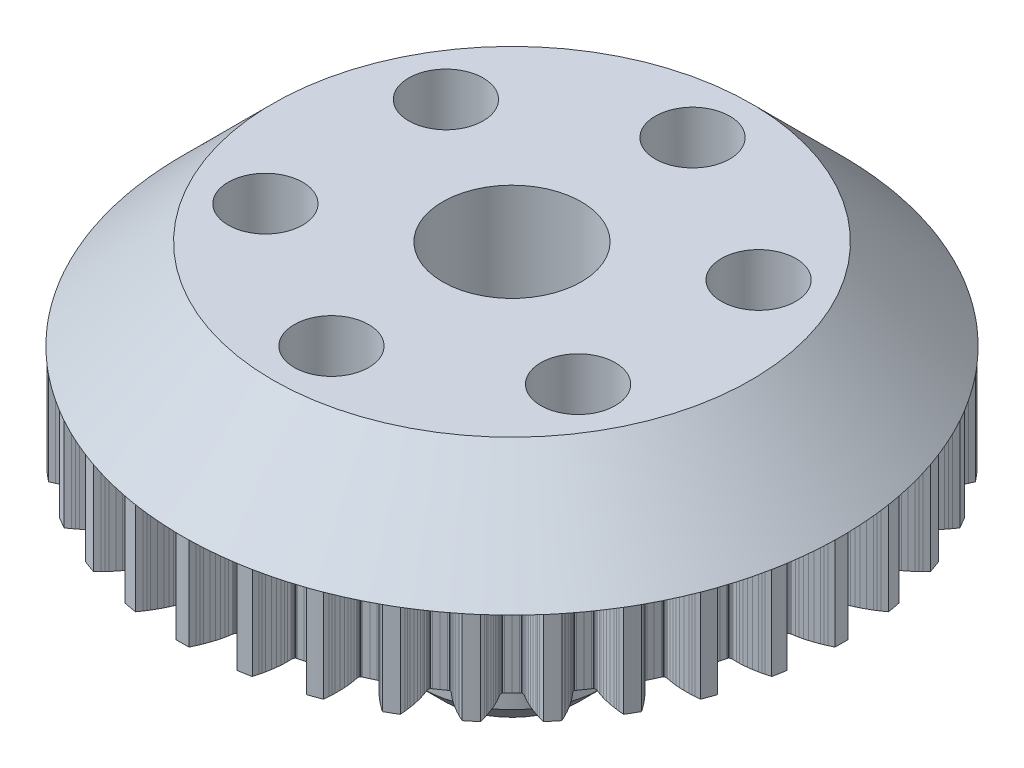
SolidWorks part; units mm, degrees
ref_plane "Front Plane" through (0, 0, 0) normal (0, 0, 1) x (1, 0, 0)
ref_plane "Top Plane" through (0, 0, 0) normal (0, 1, 0) x (1, 0, 0)
ref_plane "Right Plane" through (0, 0, 0) normal (1, 0, 0) x (0, 0, -1)
sketch "Sketch2" plane through (0, 0, 0) normal (0, 1, 0) x (1, 0, 0)
  line L632 (14.2382, 2.1155) -> (14.1321, 2.046)
  line L633 (14.1321, 2.046) -> (14.0302, 1.9822)
  line L634 (14.0302, 1.9822) -> (13.8362, 1.869)
  line L635 (13.8362, 1.869) -> (13.6574, 1.7744)
  line L636 (13.6574, 1.7744) -> (13.4969, 1.698)
  line L637 (13.4969, 1.698) -> (13.3538, 1.637)
  line L638 (13.3538, 1.637) -> (13.2277, 1.5894)
  line L639 (13.2277, 1.5894) -> (13.0788, 1.5394)
  line L640 (13.0788, 1.5394) -> (13.0417, 1.5232)
  line L641 (13.0417, 1.5232) -> (13.011, 1.5062)
  line L642 (13.011, 1.5062) -> (12.9867, 1.4887)
  line L643 (12.9867, 1.4887) -> (12.9688, 1.471)
  line L644 (12.9688, 1.471) -> (12.9574, 1.4533)
  line L645 (12.9574, 1.4533) -> (12.9524, 1.4359)
  line L646 (12.9524, 1.4359) -> (12.9583, 1.3725)
  line L647 (12.9583, 1.3725) -> (12.9811, 1.1357)
  line L648 (12.9811, 1.1357) -> (12.9998, 0.8985)
  line L649 (12.9998, 0.8985) -> (13.005, 0.8351)
  line L650 (13.005, 0.8351) -> (13.0129, 0.8188)
  line L651 (13.0129, 0.8188) -> (13.0272, 0.8034)
  line L652 (13.0272, 0.8034) -> (13.0479, 0.789)
  line L653 (13.0479, 0.789) -> (13.0749, 0.776)
  line L654 (13.0749, 0.776) -> (13.108, 0.7646)
  line L655 (13.108, 0.7646) -> (13.1474, 0.7551)
  line L656 (13.1474, 0.7551) -> (13.3028, 0.7317)
  line L657 (13.3028, 0.7317) -> (13.4352, 0.7067)
  line L658 (13.4352, 0.7067) -> (13.5867, 0.6715)
  line L659 (13.5867, 0.6715) -> (13.7581, 0.6241)
  line L660 (13.7581, 0.6241) -> (13.9505, 0.5621)
  line L662 (14.1613, 0.4843) -> (14.2727, 0.4391)
  line L663 (14.2727, 0.4391) -> (14.3893, 0.389)
  line L664 (14.3893, 0.389) -> (14.6039, 0.2893)
  line L665 (14.6039, -0.2893) -> (14.3893, -0.389)
  line L666 (14.3893, -0.389) -> (14.2727, -0.4391)
  line L667 (14.2727, -0.4391) -> (14.1613, -0.4843)
  line L668 (14.1613, -0.4843) -> (13.9505, -0.5621)
  line L669 (13.9505, -0.5621) -> (13.7581, -0.6241)
  line L670 (13.7581, -0.6241) -> (13.5867, -0.6715)
  line L671 (13.5867, -0.6715) -> (13.4352, -0.7067)
  line L672 (13.4352, -0.7067) -> (13.3028, -0.7317)
  line L673 (13.3028, -0.7317) -> (13.1474, -0.7551)
  line L674 (13.1474, -0.7551) -> (13.108, -0.7646)
  line L675 (13.108, -0.7646) -> (13.0749, -0.776)
  line L676 (13.0749, -0.776) -> (13.0479, -0.789)
  line L677 (13.0479, -0.789) -> (13.0272, -0.8034)
  line L678 (13.0272, -0.8034) -> (13.0129, -0.8188)
  line L679 (13.0129, -0.8188) -> (13.005, -0.8351)
  line L680 (13.005, -0.8351) -> (12.9998, -0.8985)
  line L681 (12.9998, -0.8985) -> (12.9811, -1.1357)
  line L682 (12.9811, -1.1357) -> (12.9583, -1.3725)
  line L683 (12.9583, -1.3725) -> (12.9524, -1.4359)
  line L684 (12.9524, -1.4359) -> (12.9574, -1.4533)
  line L685 (12.9574, -1.4533) -> (12.9688, -1.471)
  line L686 (12.9688, -1.471) -> (12.9867, -1.4887)
  line L687 (12.9867, -1.4887) -> (13.011, -1.5062)
  line L688 (13.011, -1.5062) -> (13.0417, -1.5232)
  line L689 (13.0417, -1.5232) -> (13.0788, -1.5394)
  line L690 (13.0788, -1.5394) -> (13.2277, -1.5894)
  line L691 (13.2277, -1.5894) -> (13.3538, -1.637)
  line L692 (13.3538, -1.637) -> (13.4969, -1.698)
  line L693 (13.4969, -1.698) -> (13.6574, -1.7744)
  line L694 (13.6574, -1.7744) -> (13.8362, -1.869)
  line L695 (13.8362, -1.869) -> (14.0302, -1.9822)
  line L696 (14.0302, -1.9822) -> (14.1321, -2.046)
  line L697 (14.1321, -2.046) -> (14.2382, -2.1155)
  line L698 (14.2382, -2.1155) -> (14.4322, -2.2511)
  line L699 (14.3318, -2.8208) -> (14.1031, -2.8818)
  line L700 (14.1031, -2.8818) -> (13.9796, -2.9109)
  line L701 (13.9796, -2.9109) -> (13.862, -2.936)
  line L702 (13.862, -2.936) -> (13.641, -2.976)
  line L703 (13.641, -2.976) -> (13.4407, -3.0037)
  line L704 (13.4407, -3.0037) -> (13.2637, -3.0206)
  line L705 (13.2637, -3.0206) -> (13.1084, -3.029)
  line L706 (13.1084, -3.029) -> (12.9736, -3.0306)
  line L707 (12.9736, -3.0306) -> (12.8166, -3.0266)
  line L708 (12.8166, -3.0266) -> (12.7761, -3.0292)
  line L709 (12.7761, -3.0292) -> (12.7415, -3.0347)
  line L710 (12.7415, -3.0347) -> (12.7127, -3.0428)
  line L711 (12.7127, -3.0428) -> (12.6898, -3.0534)
  line L712 (12.6898, -3.0534) -> (12.6731, -3.0661)
  line L713 (12.6731, -3.0661) -> (12.6624, -3.0807)
  line L714 (12.6624, -3.0807) -> (12.6462, -3.1422)
  line L715 (12.6462, -3.1422) -> (12.5867, -3.3726)
  line L716 (12.5867, -3.3726) -> (12.5231, -3.6019)
  line L717 (12.5231, -3.6019) -> (12.5063, -3.6632)
  line L718 (12.5063, -3.6632) -> (12.5082, -3.6812)
  line L719 (12.5082, -3.6812) -> (12.5164, -3.7006)
  line L720 (12.5164, -3.7006) -> (12.5309, -3.7212)
  line L721 (12.5309, -3.7212) -> (12.5518, -3.7426)
  line L722 (12.5518, -3.7426) -> (12.5791, -3.7647)
  line L723 (12.5791, -3.7647) -> (12.6128, -3.7872)
  line L724 (12.6128, -3.7872) -> (12.7508, -3.8623)
  line L725 (12.7508, -3.8623) -> (12.8667, -3.931)
  line L726 (12.8667, -3.931) -> (12.997, -4.0159)
  line L727 (12.997, -4.0159) -> (13.1418, -4.1191)
  line L728 (13.1418, -4.1191) -> (13.3015, -4.2432)
  line L729 (13.3015, -4.2432) -> (13.4729, -4.3884)
  line L730 (13.4729, -4.3884) -> (13.5621, -4.4689)
  line L731 (13.5621, -4.4689) -> (13.6545, -4.5558)
  line L732 (13.6545, -4.5558) -> (13.8221, -4.723)
  line L733 (13.6242, -5.2666) -> (13.3884, -5.287)
  line L734 (13.3884, -5.287) -> (13.2618, -5.2942)
  line L735 (13.2618, -5.2942) -> (13.1416, -5.2985)
  line L736 (13.1416, -5.2985) -> (12.917, -5.2995)
  line L737 (12.917, -5.2995) -> (12.7149, -5.292)
  line L738 (12.7149, -5.292) -> (12.5376, -5.2779)
  line L739 (12.5376, -5.2779) -> (12.3833, -5.2592)
  line L740 (12.3833, -5.2592) -> (12.2503, -5.2374)
  line L741 (12.2503, -5.2374) -> (12.0963, -5.2062)
  line L742 (12.0963, -5.2062) -> (12.056, -5.2017)
  line L743 (12.056, -5.2017) -> (12.0209, -5.2011)
  line L744 (12.0209, -5.2011) -> (11.9911, -5.2041)
  line L745 (11.9911, -5.2041) -> (11.9668, -5.2105)
  line L746 (11.9668, -5.2105) -> (11.9481, -5.2201)
  line L747 (11.9481, -5.2201) -> (11.9351, -5.2327)
  line L748 (11.9351, -5.2327) -> (11.9085, -5.2905)
  line L749 (11.9085, -5.2905) -> (11.8099, -5.507)
  line L750 (11.8099, -5.507) -> (11.7074, -5.7218)
  line L751 (11.7074, -5.7218) -> (11.6802, -5.7793)
  line L752 (11.6802, -5.7793) -> (11.679, -5.7973)
  line L753 (11.679, -5.7973) -> (11.6836, -5.8179)
  line L754 (11.6836, -5.8179) -> (11.6943, -5.8406)
  line L755 (11.6943, -5.8406) -> (11.7112, -5.8654)
  line L756 (11.7112, -5.8654) -> (11.7342, -5.8918)
  line L757 (11.7342, -5.8918) -> (11.7636, -5.9198)
  line L758 (11.7636, -5.9198) -> (11.8864, -6.0177)
  line L759 (11.8864, -6.0177) -> (11.9886, -6.1056)
  line L760 (11.9886, -6.1056) -> (12.1022, -6.2118)
  line L761 (12.1022, -6.2118) -> (12.2269, -6.3385)
  line L762 (12.2269, -6.3385) -> (12.3626, -6.4885)
  line L763 (12.3626, -6.4885) -> (12.5061, -6.6612)
  line L764 (12.5061, -6.6612) -> (12.5801, -6.7561)
  line L765 (12.5801, -6.7561) -> (12.656, -6.8577)
  line L766 (12.656, -6.8577) -> (12.7919, -7.0514)
  line L767 (12.5027, -7.5524) -> (12.2669, -7.5315)
  line L768 (12.2669, -7.5315) -> (12.141, -7.5166)
  line L769 (12.141, -7.5166) -> (12.0219, -7.5)
  line L770 (12.0219, -7.5) -> (11.8005, -7.462)
  line L771 (11.8005, -7.462) -> (11.6028, -7.4195)
  line L772 (11.6028, -7.4195) -> (11.4307, -7.3749)
  line L773 (11.4307, -7.3749) -> (11.2819, -7.3297)
  line L774 (11.2819, -7.3297) -> (11.1547, -7.2851)
  line L775 (11.1547, -7.2851) -> (11.0085, -7.2276)
  line L776 (11.0085, -7.2276) -> (10.9696, -7.2162)
  line L777 (10.9696, -7.2162) -> (10.9351, -7.2095)
  line L778 (10.9351, -7.2095) -> (10.9053, -7.2073)
  line L779 (10.9053, -7.2073) -> (10.8802, -7.2094)
  line L780 (10.8802, -7.2094) -> (10.8601, -7.2156)
  line L781 (10.8601, -7.2156) -> (10.8451, -7.2257)
  line L782 (10.8451, -7.2257) -> (10.8089, -7.278)
  line L783 (10.8089, -7.278) -> (10.6742, -7.4741)
  line L784 (10.6742, -7.4741) -> (10.5359, -7.6678)
  line L785 (10.5359, -7.6678) -> (10.4992, -7.7197)
  line L786 (10.4992, -7.7197) -> (10.4948, -7.7373)
  line L787 (10.4948, -7.7373) -> (10.4959, -7.7583)
  line L788 (10.4959, -7.7583) -> (10.5025, -7.7826)
  line L789 (10.5025, -7.7826) -> (10.5147, -7.8099)
  line L790 (10.5147, -7.8099) -> (10.5328, -7.84)
  line L791 (10.5328, -7.84) -> (10.5569, -7.8726)
  line L792 (10.5569, -7.8726) -> (10.6608, -7.9904)
  line L793 (10.6608, -7.9904) -> (10.7463, -8.0946)
  line L794 (10.7463, -8.0946) -> (10.8397, -8.2189)
  line L795 (10.8397, -8.2189) -> (10.9405, -8.3654)
  line L796 (10.9405, -8.3654) -> (11.048, -8.5367)
  line L797 (11.048, -8.5367) -> (11.1594, -8.7317)
  line L798 (11.1594, -8.7317) -> (11.2158, -8.8379)
  line L799 (11.2158, -8.8379) -> (11.2729, -8.9512)
  line L800 (11.2729, -8.9512) -> (11.3731, -9.1656)
  line L801 (11.0013, -9.6088) -> (10.7727, -9.5473)
  line L802 (10.7727, -9.5473) -> (10.6513, -9.5107)
  line L803 (10.6513, -9.5107) -> (10.5369, -9.4736)
  line L804 (10.5369, -9.4736) -> (10.3254, -9.3978)
  line L805 (10.3254, -9.3978) -> (10.1381, -9.3216)
  line L806 (10.1381, -9.3216) -> (9.9764, -9.2478)
  line L807 (9.9764, -9.2478) -> (9.8377, -9.1774)
  line L808 (9.8377, -9.1774) -> (9.7202, -9.1114)
  line L809 (9.7202, -9.1114) -> (9.5862, -9.0294)
  line L810 (9.5862, -9.0294) -> (9.5499, -9.0114)
  line L811 (9.5499, -9.0114) -> (9.5171, -8.9988)
  line L812 (9.5171, -8.9988) -> (9.4881, -8.9915)
  line L813 (9.4881, -8.9915) -> (9.463, -8.9892)
  line L814 (9.463, -8.9892) -> (9.4421, -8.9918)
  line L815 (9.4421, -8.9918) -> (9.4256, -8.9992)
  line L816 (9.4256, -8.9992) -> (9.3809, -9.0444)
  line L817 (9.3809, -9.0444) -> (9.2141, -9.2141)
  line L818 (9.2141, -9.2141) -> (9.0444, -9.3809)
  line L819 (9.0444, -9.3809) -> (8.9992, -9.4256)
  line L820 (8.9992, -9.4256) -> (8.9918, -9.4421)
  line L821 (8.9918, -9.4421) -> (8.9892, -9.463)
  line L822 (8.9892, -9.463) -> (8.9915, -9.4881)
  line L823 (8.9915, -9.4881) -> (8.9988, -9.5171)
  line L824 (8.9988, -9.5171) -> (9.0114, -9.5499)
  line L825 (9.0114, -9.5499) -> (9.0294, -9.5862)
  line L826 (9.0294, -9.5862) -> (9.1114, -9.7202)
  line L827 (9.1114, -9.7202) -> (9.1774, -9.8377)
  line L828 (9.1774, -9.8377) -> (9.2478, -9.9764)
  line L829 (9.2478, -9.9764) -> (9.3216, -10.1381)
  line L830 (9.3216, -10.1381) -> (9.3978, -10.3254)
  line L831 (9.3978, -10.3254) -> (9.4736, -10.5369)
  line L832 (9.4736, -10.5369) -> (9.5107, -10.6513)
  line L833 (9.5107, -10.6513) -> (9.5473, -10.7727)
  line L834 (9.5473, -10.7727) -> (9.6088, -11.0013)
  line L835 (9.1656, -11.3731) -> (8.9512, -11.2729)
  line L836 (8.9512, -11.2729) -> (8.8379, -11.2158)
  line L837 (8.8379, -11.2158) -> (8.7317, -11.1594)
  line L838 (8.7317, -11.1594) -> (8.5367, -11.048)
  line L839 (8.5367, -11.048) -> (8.3654, -10.9405)
  line L840 (8.3654, -10.9405) -> (8.2189, -10.8397)
  line L841 (8.2189, -10.8397) -> (8.0946, -10.7463)
  line L842 (8.0946, -10.7463) -> (7.9904, -10.6608)
  line L843 (7.9904, -10.6608) -> (7.8726, -10.5569)
  line L844 (7.8726, -10.5569) -> (7.84, -10.5328)
  line L845 (7.84, -10.5328) -> (7.8099, -10.5147)
  line L846 (7.8099, -10.5147) -> (7.7826, -10.5025)
  line L847 (7.7826, -10.5025) -> (7.7583, -10.4959)
  line L848 (7.7583, -10.4959) -> (7.7373, -10.4948)
  line L849 (7.7373, -10.4948) -> (7.7197, -10.4992)
  line L850 (7.7197, -10.4992) -> (7.6678, -10.5359)
  line L851 (7.6678, -10.5359) -> (7.4741, -10.6742)
  line L852 (7.4741, -10.6742) -> (7.278, -10.8089)
  line L853 (7.278, -10.8089) -> (7.2257, -10.8451)
  line L854 (7.2257, -10.8451) -> (7.2156, -10.8601)
  line L855 (7.2156, -10.8601) -> (7.2094, -10.8802)
  line L856 (7.2094, -10.8802) -> (7.2073, -10.9053)
  line L857 (7.2073, -10.9053) -> (7.2095, -10.9351)
  line L858 (7.2095, -10.9351) -> (7.2162, -10.9696)
  line L859 (7.2162, -10.9696) -> (7.2276, -11.0085)
  line L860 (7.2276, -11.0085) -> (7.2851, -11.1547)
  line L861 (7.2851, -11.1547) -> (7.3297, -11.2819)
  line L862 (7.3297, -11.2819) -> (7.3749, -11.4307)
  line L863 (7.3749, -11.4307) -> (7.4195, -11.6028)
  line L864 (7.4195, -11.6028) -> (7.462, -11.8005)
  line L865 (7.462, -11.8005) -> (7.5, -12.0219)
  line L866 (7.5, -12.0219) -> (7.5166, -12.141)
  line L867 (7.5166, -12.141) -> (7.5315, -12.2669)
  line L868 (7.5315, -12.2669) -> (7.5524, -12.5027)
  line L869 (7.0514, -12.7919) -> (6.8577, -12.656)
  line L870 (6.8577, -12.656) -> (6.7561, -12.5801)
  line L871 (6.7561, -12.5801) -> (6.6612, -12.5061)
  line L872 (6.6612, -12.5061) -> (6.4885, -12.3626)
  line L873 (6.4885, -12.3626) -> (6.3385, -12.2269)
  line L874 (6.3385, -12.2269) -> (6.2118, -12.1022)
  line L875 (6.2118, -12.1022) -> (6.1056, -11.9886)
  line L876 (6.1056, -11.9886) -> (6.0177, -11.8864)
  line L877 (6.0177, -11.8864) -> (5.9198, -11.7636)
  line L878 (5.9198, -11.7636) -> (5.8918, -11.7342)
  line L879 (5.8918, -11.7342) -> (5.8654, -11.7112)
  line L880 (5.8654, -11.7112) -> (5.8406, -11.6943)
  line L881 (5.8406, -11.6943) -> (5.8179, -11.6836)
  line L882 (5.8179, -11.6836) -> (5.7973, -11.679)
  line L883 (5.7973, -11.679) -> (5.7793, -11.6802)
  line L884 (5.7793, -11.6802) -> (5.7218, -11.7074)
  line L885 (5.7218, -11.7074) -> (5.507, -11.8099)
  line L886 (5.507, -11.8099) -> (5.2905, -11.9085)
  line L887 (5.2905, -11.9085) -> (5.2327, -11.9351)
  line L888 (5.2327, -11.9351) -> (5.2201, -11.9481)
  line L889 (5.2201, -11.9481) -> (5.2105, -11.9668)
  line L890 (5.2105, -11.9668) -> (5.2041, -11.9911)
  line L891 (5.2041, -11.9911) -> (5.2011, -12.0209)
  line L892 (5.2011, -12.0209) -> (5.2017, -12.056)
  line L893 (5.2017, -12.056) -> (5.2062, -12.0963)
  line L894 (5.2062, -12.0963) -> (5.2374, -12.2503)
  line L895 (5.2374, -12.2503) -> (5.2592, -12.3833)
  line L896 (5.2592, -12.3833) -> (5.2779, -12.5376)
  line L897 (5.2779, -12.5376) -> (5.292, -12.7149)
  line L898 (5.292, -12.7149) -> (5.2995, -12.917)
  line L899 (5.2995, -12.917) -> (5.2985, -13.1416)
  line L900 (5.2985, -13.1416) -> (5.2942, -13.2618)
  line L901 (5.2942, -13.2618) -> (5.287, -13.3884)
  line L902 (5.287, -13.3884) -> (5.2666, -13.6242)
  line L903 (4.723, -13.8221) -> (4.5558, -13.6545)
  line L904 (4.5558, -13.6545) -> (4.4689, -13.5621)
  line L905 (4.4689, -13.5621) -> (4.3884, -13.4729)
  line L906 (4.3884, -13.4729) -> (4.2432, -13.3015)
  line L907 (4.2432, -13.3015) -> (4.1191, -13.1418)
  line L908 (4.1191, -13.1418) -> (4.0159, -12.997)
  line L909 (4.0159, -12.997) -> (3.931, -12.8667)
  line L910 (3.931, -12.8667) -> (3.8623, -12.7508)
  line L911 (3.8623, -12.7508) -> (3.7872, -12.6128)
  line L912 (3.7872, -12.6128) -> (3.7647, -12.5791)
  line L913 (3.7647, -12.5791) -> (3.7426, -12.5518)
  line L914 (3.7426, -12.5518) -> (3.7212, -12.5309)
  line L915 (3.7212, -12.5309) -> (3.7006, -12.5164)
  line L916 (3.7006, -12.5164) -> (3.6812, -12.5082)
  line L917 (3.6812, -12.5082) -> (3.6632, -12.5063)
  line L918 (3.6632, -12.5063) -> (3.6019, -12.5231)
  line L919 (3.6019, -12.5231) -> (3.3726, -12.5867)
  line L920 (3.3726, -12.5867) -> (3.1422, -12.6462)
  line L921 (3.1422, -12.6462) -> (3.0807, -12.6624)
  line L922 (3.0807, -12.6624) -> (3.0661, -12.6731)
  line L923 (3.0661, -12.6731) -> (3.0534, -12.6898)
  line L924 (3.0534, -12.6898) -> (3.0428, -12.7127)
  line L925 (3.0428, -12.7127) -> (3.0347, -12.7415)
  line L926 (3.0347, -12.7415) -> (3.0292, -12.7761)
  line L927 (3.0292, -12.7761) -> (3.0266, -12.8166)
  line L928 (3.0266, -12.8166) -> (3.0306, -12.9736)
  line L929 (3.0306, -12.9736) -> (3.029, -13.1084)
  line L930 (3.029, -13.1084) -> (3.0206, -13.2637)
  line L931 (3.0206, -13.2637) -> (3.0037, -13.4407)
  line L932 (3.0037, -13.4407) -> (2.976, -13.641)
  line L933 (2.976, -13.641) -> (2.936, -13.862)
  line L934 (2.936, -13.862) -> (2.9109, -13.9796)
  line L935 (2.9109, -13.9796) -> (2.8818, -14.1031)
  line L936 (2.8818, -14.1031) -> (2.8208, -14.3318)
  line L937 (2.2511, -14.4322) -> (2.1155, -14.2382)
  line L938 (2.1155, -14.2382) -> (2.046, -14.1321)
  line L939 (2.046, -14.1321) -> (1.9822, -14.0302)
  line L940 (1.9822, -14.0302) -> (1.869, -13.8362)
  line L941 (1.869, -13.8362) -> (1.7744, -13.6574)
  line L942 (1.7744, -13.6574) -> (1.698, -13.4969)
  line L943 (1.698, -13.4969) -> (1.637, -13.3538)
  line L944 (1.637, -13.3538) -> (1.5894, -13.2277)
  line L945 (1.5894, -13.2277) -> (1.5394, -13.0788)
  line L946 (1.5394, -13.0788) -> (1.5232, -13.0417)
  line L947 (1.5232, -13.0417) -> (1.5062, -13.011)
  line L948 (1.5062, -13.011) -> (1.4887, -12.9867)
  line L949 (1.4887, -12.9867) -> (1.471, -12.9688)
  line L950 (1.471, -12.9688) -> (1.4533, -12.9574)
  line L951 (1.4533, -12.9574) -> (1.4359, -12.9524)
  line L952 (1.4359, -12.9524) -> (1.3725, -12.9583)
  line L953 (1.3725, -12.9583) -> (1.1357, -12.9811)
  line L954 (1.1357, -12.9811) -> (0.8985, -12.9998)
  line L955 (0.8985, -12.9998) -> (0.8351, -13.005)
  line L956 (0.8351, -13.005) -> (0.8188, -13.0129)
  line L957 (0.8188, -13.0129) -> (0.8034, -13.0272)
  line L958 (0.8034, -13.0272) -> (0.789, -13.0479)
  line L959 (0.789, -13.0479) -> (0.776, -13.0749)
  line L960 (0.776, -13.0749) -> (0.7646, -13.108)
  line L961 (0.7646, -13.108) -> (0.7551, -13.1474)
  line L962 (0.7551, -13.1474) -> (0.7317, -13.3028)
  line L963 (0.7317, -13.3028) -> (0.7067, -13.4352)
  line L964 (0.7067, -13.4352) -> (0.6715, -13.5867)
  line L965 (0.6715, -13.5867) -> (0.6241, -13.7581)
  line L966 (0.6241, -13.7581) -> (0.5621, -13.9505)
  line L967 (0.5621, -13.9505) -> (0.4843, -14.1613)
  line L968 (0.4843, -14.1613) -> (0.4391, -14.2727)
  line L969 (0.4391, -14.2727) -> (0.389, -14.3893)
  line L970 (0.389, -14.3893) -> (0.2893, -14.6039)
  line L971 (-0.2893, -14.6039) -> (-0.389, -14.3893)
  line L972 (-0.389, -14.3893) -> (-0.4391, -14.2727)
  line L973 (-0.4391, -14.2727) -> (-0.4843, -14.1613)
  line L974 (-0.4843, -14.1613) -> (-0.5621, -13.9505)
  line L975 (-0.5621, -13.9505) -> (-0.6241, -13.7581)
  line L976 (-0.6241, -13.7581) -> (-0.6715, -13.5867)
  line L977 (-0.6715, -13.5867) -> (-0.7067, -13.4352)
  line L978 (-0.7067, -13.4352) -> (-0.7317, -13.3028)
  line L979 (-0.7317, -13.3028) -> (-0.7551, -13.1474)
  line L980 (-0.7551, -13.1474) -> (-0.7646, -13.108)
  line L981 (-0.7646, -13.108) -> (-0.776, -13.0749)
  line L982 (-0.776, -13.0749) -> (-0.789, -13.0479)
  line L983 (-0.789, -13.0479) -> (-0.8034, -13.0272)
  line L984 (-0.8034, -13.0272) -> (-0.8188, -13.0129)
  line L985 (-0.8188, -13.0129) -> (-0.8351, -13.005)
  line L986 (-0.8351, -13.005) -> (-0.8985, -12.9998)
  line L987 (-0.8985, -12.9998) -> (-1.1357, -12.9811)
  line L988 (-1.1357, -12.9811) -> (-1.3725, -12.9583)
  line L989 (-1.3725, -12.9583) -> (-1.4359, -12.9524)
  line L990 (-1.4359, -12.9524) -> (-1.4533, -12.9574)
  line L991 (-1.4533, -12.9574) -> (-1.471, -12.9688)
  line L992 (-1.471, -12.9688) -> (-1.4887, -12.9867)
  line L993 (-1.4887, -12.9867) -> (-1.5062, -13.011)
  line L994 (-1.5062, -13.011) -> (-1.5232, -13.0417)
  line L995 (-1.5232, -13.0417) -> (-1.5394, -13.0788)
  line L996 (-1.5394, -13.0788) -> (-1.5894, -13.2277)
  line L997 (-1.5894, -13.2277) -> (-1.637, -13.3538)
  line L998 (-1.637, -13.3538) -> (-1.698, -13.4969)
  line L999 (-1.698, -13.4969) -> (-1.7744, -13.6574)
  line L1000 (-1.7744, -13.6574) -> (-1.869, -13.8362)
  line L1001 (-1.869, -13.8362) -> (-1.9822, -14.0302)
  line L1002 (-1.9822, -14.0302) -> (-2.046, -14.1321)
  line L1003 (-2.046, -14.1321) -> (-2.1155, -14.2382)
  line L1004 (-2.1155, -14.2382) -> (-2.2511, -14.4322)
  line L1005 (-2.8208, -14.3318) -> (-2.8818, -14.1031)
  line L1006 (-2.8818, -14.1031) -> (-2.9109, -13.9796)
  line L1007 (-2.9109, -13.9796) -> (-2.936, -13.862)
  line L1008 (-2.936, -13.862) -> (-2.976, -13.641)
  line L1009 (-2.976, -13.641) -> (-3.0037, -13.4407)
  line L1010 (-3.0037, -13.4407) -> (-3.0206, -13.2637)
  line L1011 (-3.0206, -13.2637) -> (-3.029, -13.1084)
  line L1012 (-3.029, -13.1084) -> (-3.0306, -12.9736)
  line L1013 (-3.0306, -12.9736) -> (-3.0266, -12.8166)
  line L1014 (-3.0266, -12.8166) -> (-3.0292, -12.7761)
  line L1015 (-3.0292, -12.7761) -> (-3.0347, -12.7415)
  line L1016 (-3.0347, -12.7415) -> (-3.0428, -12.7127)
  line L1017 (-3.0428, -12.7127) -> (-3.0534, -12.6898)
  line L1018 (-3.0534, -12.6898) -> (-3.0661, -12.6731)
  line L1019 (-3.0661, -12.6731) -> (-3.0807, -12.6624)
  line L1020 (-3.0807, -12.6624) -> (-3.1422, -12.6462)
  line L1021 (-3.1422, -12.6462) -> (-3.3726, -12.5867)
  line L1022 (-3.3726, -12.5867) -> (-3.6019, -12.5231)
  line L1023 (-3.6019, -12.5231) -> (-3.6632, -12.5063)
  line L1024 (-3.6632, -12.5063) -> (-3.6812, -12.5082)
  line L1025 (-3.6812, -12.5082) -> (-3.7006, -12.5164)
  line L1026 (-3.7006, -12.5164) -> (-3.7212, -12.5309)
  line L1027 (-3.7212, -12.5309) -> (-3.7426, -12.5518)
  line L1028 (-3.7426, -12.5518) -> (-3.7647, -12.5791)
  line L1029 (-3.7647, -12.5791) -> (-3.7872, -12.6128)
  line L1030 (-3.7872, -12.6128) -> (-3.8623, -12.7508)
  line L1031 (-3.8623, -12.7508) -> (-3.931, -12.8667)
  line L1032 (-3.931, -12.8667) -> (-4.0159, -12.997)
  line L1033 (-4.0159, -12.997) -> (-4.1191, -13.1418)
  line L1034 (-4.1191, -13.1418) -> (-4.2432, -13.3015)
  line L1035 (-4.2432, -13.3015) -> (-4.3884, -13.4729)
  line L1036 (-4.3884, -13.4729) -> (-4.4689, -13.5621)
  line L1037 (-4.4689, -13.5621) -> (-4.5558, -13.6545)
  line L1038 (-4.5558, -13.6545) -> (-4.723, -13.8221)
  line L1039 (-5.2666, -13.6242) -> (-5.287, -13.3884)
  line L1040 (-5.287, -13.3884) -> (-5.2942, -13.2618)
  line L1041 (-5.2942, -13.2618) -> (-5.2985, -13.1416)
  line L1042 (-5.2985, -13.1416) -> (-5.2995, -12.917)
  line L1043 (-5.2995, -12.917) -> (-5.292, -12.7149)
  line L1044 (-5.292, -12.7149) -> (-5.2779, -12.5376)
  line L1045 (-5.2779, -12.5376) -> (-5.2592, -12.3833)
  line L1046 (-5.2592, -12.3833) -> (-5.2374, -12.2503)
  line L1047 (-5.2374, -12.2503) -> (-5.2062, -12.0963)
  line L1048 (-5.2062, -12.0963) -> (-5.2017, -12.056)
  line L1049 (-5.2017, -12.056) -> (-5.2011, -12.0209)
  line L1050 (-5.2011, -12.0209) -> (-5.2041, -11.9911)
  line L1051 (-5.2041, -11.9911) -> (-5.2105, -11.9668)
  line L1052 (-5.2105, -11.9668) -> (-5.2201, -11.9481)
  line L1053 (-5.2201, -11.9481) -> (-5.2327, -11.9351)
  line L1054 (-5.2327, -11.9351) -> (-5.2905, -11.9085)
  line L1055 (-5.2905, -11.9085) -> (-5.507, -11.8099)
  line L1056 (-5.507, -11.8099) -> (-5.7218, -11.7074)
  line L1057 (-5.7218, -11.7074) -> (-5.7793, -11.6802)
  line L1058 (-5.7793, -11.6802) -> (-5.7973, -11.679)
  line L1059 (-5.7973, -11.679) -> (-5.8179, -11.6836)
  line L1060 (-5.8179, -11.6836) -> (-5.8406, -11.6943)
  line L1061 (-5.8406, -11.6943) -> (-5.8654, -11.7112)
  line L1062 (-5.8654, -11.7112) -> (-5.8918, -11.7342)
  line L1063 (-5.8918, -11.7342) -> (-5.9198, -11.7636)
  line L1064 (-5.9198, -11.7636) -> (-6.0177, -11.8864)
  line L1065 (-6.0177, -11.8864) -> (-6.1056, -11.9886)
  line L1066 (-6.1056, -11.9886) -> (-6.2118, -12.1022)
  line L1067 (-6.2118, -12.1022) -> (-6.3385, -12.2269)
  line L1068 (-6.3385, -12.2269) -> (-6.4885, -12.3626)
  line L1069 (-6.4885, -12.3626) -> (-6.6612, -12.5061)
  line L1070 (-6.6612, -12.5061) -> (-6.7561, -12.5801)
  line L1071 (-6.7561, -12.5801) -> (-6.8577, -12.656)
  line L1072 (-6.8577, -12.656) -> (-7.0514, -12.7919)
  line L1073 (-7.5524, -12.5027) -> (-7.5315, -12.2669)
  line L1074 (-7.5315, -12.2669) -> (-7.5166, -12.141)
  line L1075 (-7.5166, -12.141) -> (-7.5, -12.0219)
  line L1076 (-7.5, -12.0219) -> (-7.462, -11.8005)
  line L1077 (-7.462, -11.8005) -> (-7.4195, -11.6028)
  line L1078 (-7.4195, -11.6028) -> (-7.3749, -11.4307)
  line L1079 (-7.3749, -11.4307) -> (-7.3297, -11.2819)
  line L1080 (-7.3297, -11.2819) -> (-7.2851, -11.1547)
  line L1081 (-7.2851, -11.1547) -> (-7.2276, -11.0085)
  line L1082 (-7.2276, -11.0085) -> (-7.2162, -10.9696)
  line L1083 (-7.2162, -10.9696) -> (-7.2095, -10.9351)
  line L1084 (-7.2095, -10.9351) -> (-7.2073, -10.9053)
  line L1085 (-7.2073, -10.9053) -> (-7.2094, -10.8802)
  line L1086 (-7.2094, -10.8802) -> (-7.2156, -10.8601)
  line L1087 (-7.2156, -10.8601) -> (-7.2257, -10.8451)
  line L1088 (-7.2257, -10.8451) -> (-7.278, -10.8089)
  line L1089 (-7.278, -10.8089) -> (-7.4741, -10.6742)
  line L1090 (-7.4741, -10.6742) -> (-7.6678, -10.5359)
  line L1091 (-7.6678, -10.5359) -> (-7.7197, -10.4992)
  line L1092 (-7.7197, -10.4992) -> (-7.7373, -10.4948)
  line L1093 (-7.7373, -10.4948) -> (-7.7583, -10.4959)
  line L1094 (-7.7583, -10.4959) -> (-7.7826, -10.5025)
  line L1095 (-7.7826, -10.5025) -> (-7.8099, -10.5147)
  line L1096 (-7.8099, -10.5147) -> (-7.84, -10.5328)
  line L1097 (-7.84, -10.5328) -> (-7.8726, -10.5569)
  line L1098 (-7.8726, -10.5569) -> (-7.9904, -10.6608)
  line L1099 (-7.9904, -10.6608) -> (-8.0946, -10.7463)
  line L1100 (-8.0946, -10.7463) -> (-8.2189, -10.8397)
  line L1101 (-8.2189, -10.8397) -> (-8.3654, -10.9405)
  line L1102 (-8.3654, -10.9405) -> (-8.5367, -11.048)
  line L1103 (-8.5367, -11.048) -> (-8.7317, -11.1594)
  line L1104 (-8.7317, -11.1594) -> (-8.8379, -11.2158)
  line L1105 (-8.8379, -11.2158) -> (-8.9512, -11.2729)
  line L1106 (-8.9512, -11.2729) -> (-9.1656, -11.3731)
  line L1107 (-9.6088, -11.0013) -> (-9.5473, -10.7727)
  line L1108 (-9.5473, -10.7727) -> (-9.5107, -10.6513)
  line L1109 (-9.5107, -10.6513) -> (-9.4736, -10.5369)
  line L1110 (-9.4736, -10.5369) -> (-9.3978, -10.3254)
  line L1111 (-9.3978, -10.3254) -> (-9.3216, -10.1381)
  line L1112 (-9.3216, -10.1381) -> (-9.2478, -9.9764)
  line L1113 (-9.2478, -9.9764) -> (-9.1774, -9.8377)
  line L1114 (-9.1774, -9.8377) -> (-9.1114, -9.7202)
  line L1115 (-9.1114, -9.7202) -> (-9.0294, -9.5862)
  line L1116 (-9.0294, -9.5862) -> (-9.0114, -9.5499)
  line L1117 (-9.0114, -9.5499) -> (-8.9988, -9.5171)
  line L1118 (-8.9988, -9.5171) -> (-8.9915, -9.4881)
  line L1119 (-8.9915, -9.4881) -> (-8.9892, -9.463)
  line L1120 (-8.9892, -9.463) -> (-8.9918, -9.4421)
  line L1121 (-8.9918, -9.4421) -> (-8.9992, -9.4256)
  line L1122 (-8.9992, -9.4256) -> (-9.0444, -9.3809)
  line L1123 (-9.0444, -9.3809) -> (-9.2141, -9.2141)
  line L1124 (-9.2141, -9.2141) -> (-9.3809, -9.0444)
  line L1125 (-9.3809, -9.0444) -> (-9.4256, -8.9992)
  line L1126 (-9.4256, -8.9992) -> (-9.4421, -8.9918)
  line L1127 (-9.4421, -8.9918) -> (-9.463, -8.9892)
  line L1128 (-9.463, -8.9892) -> (-9.4881, -8.9915)
  line L1129 (-9.4881, -8.9915) -> (-9.5171, -8.9988)
  line L1130 (-9.5171, -8.9988) -> (-9.5499, -9.0114)
  line L1131 (-9.5499, -9.0114) -> (-9.5862, -9.0294)
  line L1132 (-9.5862, -9.0294) -> (-9.7202, -9.1114)
  line L1133 (-9.7202, -9.1114) -> (-9.8377, -9.1774)
  line L1134 (-9.8377, -9.1774) -> (-9.9764, -9.2478)
  line L1135 (-9.9764, -9.2478) -> (-10.1381, -9.3216)
  line L1136 (-10.1381, -9.3216) -> (-10.3254, -9.3978)
  line L1137 (-10.3254, -9.3978) -> (-10.5369, -9.4736)
  line L1138 (-10.5369, -9.4736) -> (-10.6513, -9.5107)
  line L1139 (-10.6513, -9.5107) -> (-10.7727, -9.5473)
  line L1140 (-10.7727, -9.5473) -> (-11.0013, -9.6088)
  line L1141 (-11.3731, -9.1656) -> (-11.2729, -8.9512)
  line L1142 (-11.2729, -8.9512) -> (-11.2158, -8.8379)
  line L1143 (-11.2158, -8.8379) -> (-11.1594, -8.7317)
  line L1144 (-11.1594, -8.7317) -> (-11.048, -8.5367)
  line L1145 (-11.048, -8.5367) -> (-10.9405, -8.3654)
  line L1146 (-10.9405, -8.3654) -> (-10.8397, -8.2189)
  line L1147 (-10.8397, -8.2189) -> (-10.7463, -8.0946)
  line L1148 (-10.7463, -8.0946) -> (-10.6608, -7.9904)
  line L1149 (-10.6608, -7.9904) -> (-10.5569, -7.8726)
  line L1150 (-10.5569, -7.8726) -> (-10.5328, -7.84)
  line L1151 (-10.5328, -7.84) -> (-10.5147, -7.8099)
  line L1152 (-10.5147, -7.8099) -> (-10.5025, -7.7826)
  line L1153 (-10.5025, -7.7826) -> (-10.4959, -7.7583)
  line L1154 (-10.4959, -7.7583) -> (-10.4948, -7.7373)
  line L1155 (-10.4948, -7.7373) -> (-10.4992, -7.7197)
  line L1156 (-10.4992, -7.7197) -> (-10.5359, -7.6678)
  line L1157 (-10.5359, -7.6678) -> (-10.6742, -7.4741)
  line L1158 (-10.6742, -7.4741) -> (-10.8089, -7.278)
  line L1159 (-10.8089, -7.278) -> (-10.8451, -7.2257)
  line L1160 (-10.8451, -7.2257) -> (-10.8601, -7.2156)
  line L1161 (-10.8601, -7.2156) -> (-10.8802, -7.2094)
  line L1162 (-10.8802, -7.2094) -> (-10.9053, -7.2073)
  line L1163 (-10.9053, -7.2073) -> (-10.9351, -7.2095)
  line L1164 (-10.9351, -7.2095) -> (-10.9696, -7.2162)
  line L1165 (-10.9696, -7.2162) -> (-11.0085, -7.2276)
  line L1166 (-11.0085, -7.2276) -> (-11.1547, -7.2851)
  line L1167 (-11.1547, -7.2851) -> (-11.2819, -7.3297)
  line L1168 (-11.2819, -7.3297) -> (-11.4307, -7.3749)
  line L1169 (-11.4307, -7.3749) -> (-11.6028, -7.4195)
  line L1170 (-11.6028, -7.4195) -> (-11.8005, -7.462)
  line L1171 (-11.8005, -7.462) -> (-12.0219, -7.5)
  line L1172 (-12.0219, -7.5) -> (-12.141, -7.5166)
  line L1173 (-12.141, -7.5166) -> (-12.2669, -7.5315)
  line L1174 (-12.2669, -7.5315) -> (-12.5027, -7.5524)
  line L1175 (-12.7919, -7.0514) -> (-12.656, -6.8577)
  line L1176 (-12.656, -6.8577) -> (-12.5801, -6.7561)
  line L1177 (-12.5801, -6.7561) -> (-12.5061, -6.6612)
  line L1178 (-12.5061, -6.6612) -> (-12.3626, -6.4885)
  line L1179 (-12.3626, -6.4885) -> (-12.2269, -6.3385)
  line L1180 (-12.2269, -6.3385) -> (-12.1022, -6.2118)
  line L1181 (-12.1022, -6.2118) -> (-11.9886, -6.1056)
  line L1182 (-11.9886, -6.1056) -> (-11.8864, -6.0177)
  line L1183 (-11.8864, -6.0177) -> (-11.7636, -5.9198)
  line L1184 (-11.7636, -5.9198) -> (-11.7342, -5.8918)
  line L1185 (-11.7342, -5.8918) -> (-11.7112, -5.8654)
  line L1186 (-11.7112, -5.8654) -> (-11.6943, -5.8406)
  line L1187 (-11.6943, -5.8406) -> (-11.6836, -5.8179)
  line L1188 (-11.6836, -5.8179) -> (-11.679, -5.7973)
  line L1189 (-11.679, -5.7973) -> (-11.6802, -5.7793)
  line L1190 (-11.6802, -5.7793) -> (-11.7074, -5.7218)
  line L1191 (-11.7074, -5.7218) -> (-11.8099, -5.507)
  line L1192 (-11.8099, -5.507) -> (-11.9085, -5.2905)
  line L1193 (-11.9085, -5.2905) -> (-11.9351, -5.2327)
  line L1194 (-11.9351, -5.2327) -> (-11.9481, -5.2201)
  line L1195 (-11.9481, -5.2201) -> (-11.9668, -5.2105)
  line L1196 (-11.9668, -5.2105) -> (-11.9911, -5.2041)
  line L1197 (-11.9911, -5.2041) -> (-12.0209, -5.2011)
  line L1198 (-12.0209, -5.2011) -> (-12.056, -5.2017)
  line L1199 (-12.056, -5.2017) -> (-12.0963, -5.2062)
  line L1200 (-12.0963, -5.2062) -> (-12.2503, -5.2374)
  line L1201 (-12.2503, -5.2374) -> (-12.3833, -5.2592)
  line L1202 (-12.3833, -5.2592) -> (-12.5376, -5.2779)
  line L1203 (-12.5376, -5.2779) -> (-12.7149, -5.292)
  line L1204 (-12.7149, -5.292) -> (-12.917, -5.2995)
  line L1205 (-12.917, -5.2995) -> (-13.1416, -5.2985)
  line L1206 (-13.1416, -5.2985) -> (-13.2618, -5.2942)
  line L1207 (-13.2618, -5.2942) -> (-13.3884, -5.287)
  line L1208 (-13.3884, -5.287) -> (-13.6242, -5.2666)
  line L1209 (-13.8221, -4.723) -> (-13.6545, -4.5558)
  line L1210 (-13.6545, -4.5558) -> (-13.5621, -4.4689)
  line L1211 (-13.5621, -4.4689) -> (-13.4729, -4.3884)
  line L1212 (-13.4729, -4.3884) -> (-13.3015, -4.2432)
  line L1213 (-13.3015, -4.2432) -> (-13.1418, -4.1191)
  line L1214 (-13.1418, -4.1191) -> (-12.997, -4.0159)
  line L1215 (-12.997, -4.0159) -> (-12.8667, -3.931)
  line L1216 (-12.8667, -3.931) -> (-12.7508, -3.8623)
  line L1217 (-12.7508, -3.8623) -> (-12.6128, -3.7872)
  line L1218 (-12.6128, -3.7872) -> (-12.5791, -3.7647)
  line L1219 (-12.5791, -3.7647) -> (-12.5518, -3.7426)
  line L1220 (-12.5518, -3.7426) -> (-12.5309, -3.7212)
  line L1221 (-12.5309, -3.7212) -> (-12.5164, -3.7006)
  line L1222 (-12.5164, -3.7006) -> (-12.5082, -3.6812)
  line L1223 (-12.5082, -3.6812) -> (-12.5063, -3.6632)
  line L1224 (-12.5063, -3.6632) -> (-12.5231, -3.6019)
  line L1225 (-12.5231, -3.6019) -> (-12.5867, -3.3726)
  line L1226 (-12.5867, -3.3726) -> (-12.6462, -3.1422)
  line L1227 (-12.6462, -3.1422) -> (-12.6624, -3.0807)
  line L1228 (-12.6624, -3.0807) -> (-12.6731, -3.0661)
  line L1229 (-12.6731, -3.0661) -> (-12.6898, -3.0534)
  line L1230 (-12.6898, -3.0534) -> (-12.7127, -3.0428)
  line L1231 (-12.7127, -3.0428) -> (-12.7415, -3.0347)
  line L1232 (-12.7415, -3.0347) -> (-12.7761, -3.0292)
  line L1233 (-12.7761, -3.0292) -> (-12.8166, -3.0266)
  line L1234 (-12.8166, -3.0266) -> (-12.9736, -3.0306)
  line L1235 (-12.9736, -3.0306) -> (-13.1084, -3.029)
  line L1236 (-13.1084, -3.029) -> (-13.2637, -3.0206)
  line L1237 (-13.2637, -3.0206) -> (-13.4407, -3.0037)
  line L1238 (-13.4407, -3.0037) -> (-13.641, -2.976)
  line L1239 (-13.641, -2.976) -> (-13.862, -2.936)
  line L1240 (-13.862, -2.936) -> (-13.9796, -2.9109)
  line L1241 (-13.9796, -2.9109) -> (-14.1031, -2.8818)
  line L1242 (-14.1031, -2.8818) -> (-14.3318, -2.8208)
  line L1243 (-14.4322, -2.2511) -> (-14.2382, -2.1155)
  line L1244 (-14.2382, -2.1155) -> (-14.1321, -2.046)
  line L1245 (-14.1321, -2.046) -> (-14.0302, -1.9822)
  line L1246 (-14.0302, -1.9822) -> (-13.8362, -1.869)
  line L1247 (-13.8362, -1.869) -> (-13.6574, -1.7744)
  line L1248 (-13.6574, -1.7744) -> (-13.4969, -1.698)
  line L1249 (-13.4969, -1.698) -> (-13.3538, -1.637)
  line L1250 (-13.3538, -1.637) -> (-13.2277, -1.5894)
  line L1251 (-13.2277, -1.5894) -> (-13.0788, -1.5394)
  line L1252 (-13.0788, -1.5394) -> (-13.0417, -1.5232)
  line L1253 (-13.0417, -1.5232) -> (-13.011, -1.5062)
  line L1254 (-13.011, -1.5062) -> (-12.9867, -1.4887)
  line L1255 (-12.9867, -1.4887) -> (-12.9688, -1.471)
  line L1256 (-12.9688, -1.471) -> (-12.9574, -1.4533)
  line L1257 (-12.9574, -1.4533) -> (-12.9524, -1.4359)
  line L1258 (-12.9524, -1.4359) -> (-12.9583, -1.3725)
  line L1259 (-12.9583, -1.3725) -> (-12.9811, -1.1357)
  line L1260 (-12.9811, -1.1357) -> (-12.9998, -0.8985)
  line L1261 (-12.9998, -0.8985) -> (-13.005, -0.8351)
  line L1262 (-13.005, -0.8351) -> (-13.0129, -0.8188)
  line L1263 (-13.0129, -0.8188) -> (-13.0272, -0.8034)
  line L1264 (-13.0272, -0.8034) -> (-13.0479, -0.789)
  line L1265 (-13.0479, -0.789) -> (-13.0749, -0.776)
  line L1266 (-13.0749, -0.776) -> (-13.108, -0.7646)
  line L1267 (-13.108, -0.7646) -> (-13.1474, -0.7551)
  line L1268 (-13.1474, -0.7551) -> (-13.3028, -0.7317)
  line L1269 (-13.3028, -0.7317) -> (-13.4352, -0.7067)
  line L1270 (-13.4352, -0.7067) -> (-13.5867, -0.6715)
  line L1271 (-13.5867, -0.6715) -> (-13.7581, -0.6241)
  line L1272 (-13.7581, -0.6241) -> (-13.9505, -0.5621)
  line L1273 (-13.9505, -0.5621) -> (-14.1613, -0.4843)
  line L1274 (-14.1613, -0.4843) -> (-14.2727, -0.4391)
  line L1275 (-14.2727, -0.4391) -> (-14.3893, -0.389)
  line L1276 (-14.3893, -0.389) -> (-14.6039, -0.2893)
  line L1277 (-14.6039, 0.2893) -> (-14.3893, 0.389)
  line L1278 (-14.3893, 0.389) -> (-14.2727, 0.4391)
  line L1279 (-14.2727, 0.4391) -> (-14.1613, 0.4843)
  line L1280 (-14.1613, 0.4843) -> (-13.9505, 0.5621)
  line L1281 (-13.9505, 0.5621) -> (-13.7581, 0.6241)
  line L1282 (-13.7581, 0.6241) -> (-13.5867, 0.6715)
  line L1283 (-13.5867, 0.6715) -> (-13.4352, 0.7067)
  line L1284 (-13.4352, 0.7067) -> (-13.3028, 0.7317)
  line L1285 (-13.3028, 0.7317) -> (-13.1474, 0.7551)
  line L1286 (-13.1474, 0.7551) -> (-13.108, 0.7646)
  line L1287 (-13.108, 0.7646) -> (-13.0749, 0.776)
  line L1288 (-13.0749, 0.776) -> (-13.0479, 0.789)
  line L1289 (-13.0479, 0.789) -> (-13.0272, 0.8034)
  line L1290 (-13.0272, 0.8034) -> (-13.0129, 0.8188)
  line L1291 (-13.0129, 0.8188) -> (-13.005, 0.8351)
  line L1292 (-13.005, 0.8351) -> (-12.9998, 0.8985)
  line L1293 (-12.9998, 0.8985) -> (-12.9811, 1.1357)
  line L1294 (-12.9811, 1.1357) -> (-12.9583, 1.3725)
  line L1295 (-12.9583, 1.3725) -> (-12.9524, 1.4359)
  line L1296 (-12.9524, 1.4359) -> (-12.9574, 1.4533)
  line L1297 (-12.9574, 1.4533) -> (-12.9688, 1.471)
  line L1298 (-12.9688, 1.471) -> (-12.9867, 1.4887)
  line L1299 (-12.9867, 1.4887) -> (-13.011, 1.5062)
  line L1300 (-13.011, 1.5062) -> (-13.0417, 1.5232)
  line L1301 (-13.0417, 1.5232) -> (-13.0788, 1.5394)
  line L1302 (-13.0788, 1.5394) -> (-13.2277, 1.5894)
  line L1303 (-13.2277, 1.5894) -> (-13.3538, 1.637)
  line L1304 (-13.3538, 1.637) -> (-13.4969, 1.698)
  line L1305 (-13.4969, 1.698) -> (-13.6574, 1.7744)
  line L1306 (-13.6574, 1.7744) -> (-13.8362, 1.869)
  line L1307 (-13.8362, 1.869) -> (-14.0302, 1.9822)
  line L1308 (-14.0302, 1.9822) -> (-14.1321, 2.046)
  line L1309 (-14.1321, 2.046) -> (-14.2382, 2.1155)
  line L1310 (-14.2382, 2.1155) -> (-14.4322, 2.2511)
  line L1311 (-14.3318, 2.8208) -> (-14.1031, 2.8818)
  line L1312 (-14.1031, 2.8818) -> (-13.9796, 2.9109)
  line L1313 (-13.9796, 2.9109) -> (-13.862, 2.936)
  line L1314 (-13.862, 2.936) -> (-13.641, 2.976)
  line L1315 (-13.641, 2.976) -> (-13.4407, 3.0037)
  line L1316 (-13.4407, 3.0037) -> (-13.2637, 3.0206)
  line L1317 (-13.2637, 3.0206) -> (-13.1084, 3.029)
  line L1318 (-13.1084, 3.029) -> (-12.9736, 3.0306)
  line L1319 (-12.9736, 3.0306) -> (-12.8166, 3.0266)
  line L1320 (-12.8166, 3.0266) -> (-12.7761, 3.0292)
  line L1321 (-12.7761, 3.0292) -> (-12.7415, 3.0347)
  line L1322 (-12.7415, 3.0347) -> (-12.7127, 3.0428)
  line L1323 (-12.7127, 3.0428) -> (-12.6898, 3.0534)
  line L1324 (-12.6898, 3.0534) -> (-12.6731, 3.0661)
  line L1325 (-12.6731, 3.0661) -> (-12.6624, 3.0807)
  line L1326 (-12.6624, 3.0807) -> (-12.6462, 3.1422)
  line L1327 (-12.6462, 3.1422) -> (-12.5867, 3.3726)
  line L1328 (-12.5867, 3.3726) -> (-12.5231, 3.6019)
  line L1329 (-12.5231, 3.6019) -> (-12.5063, 3.6632)
  line L1330 (-12.5063, 3.6632) -> (-12.5082, 3.6812)
  line L1331 (-12.5082, 3.6812) -> (-12.5164, 3.7006)
  line L1332 (-12.5164, 3.7006) -> (-12.5309, 3.7212)
  line L1333 (-12.5309, 3.7212) -> (-12.5518, 3.7426)
  line L1334 (-12.5518, 3.7426) -> (-12.5791, 3.7647)
  line L1335 (-12.5791, 3.7647) -> (-12.6128, 3.7872)
  line L1336 (-12.6128, 3.7872) -> (-12.7508, 3.8623)
  line L1337 (-12.7508, 3.8623) -> (-12.8667, 3.931)
  line L1338 (-12.8667, 3.931) -> (-12.997, 4.0159)
  line L1339 (-12.997, 4.0159) -> (-13.1418, 4.1191)
  line L1340 (-13.1418, 4.1191) -> (-13.3015, 4.2432)
  line L1341 (-13.3015, 4.2432) -> (-13.4729, 4.3884)
  line L1342 (-13.4729, 4.3884) -> (-13.5621, 4.4689)
  line L1343 (-13.5621, 4.4689) -> (-13.6545, 4.5558)
  line L1344 (-13.6545, 4.5558) -> (-13.8221, 4.723)
  line L1345 (-13.6242, 5.2666) -> (-13.3884, 5.287)
  line L1346 (-13.3884, 5.287) -> (-13.2618, 5.2942)
  line L1347 (-13.2618, 5.2942) -> (-13.1416, 5.2985)
  line L1348 (-13.1416, 5.2985) -> (-12.917, 5.2995)
  line L1349 (-12.917, 5.2995) -> (-12.7149, 5.292)
  line L1350 (-12.7149, 5.292) -> (-12.5376, 5.2779)
  line L1351 (-12.5376, 5.2779) -> (-12.3833, 5.2592)
  line L1352 (-12.3833, 5.2592) -> (-12.2503, 5.2374)
  line L1353 (-12.2503, 5.2374) -> (-12.0963, 5.2062)
  line L1354 (-12.0963, 5.2062) -> (-12.056, 5.2017)
  line L1355 (-12.056, 5.2017) -> (-12.0209, 5.2011)
  line L1356 (-12.0209, 5.2011) -> (-11.9911, 5.2041)
  line L1357 (-11.9911, 5.2041) -> (-11.9668, 5.2105)
  line L1358 (-11.9668, 5.2105) -> (-11.9481, 5.2201)
  line L1359 (-11.9481, 5.2201) -> (-11.9351, 5.2327)
  line L1360 (-11.9351, 5.2327) -> (-11.9085, 5.2905)
  line L1361 (-11.9085, 5.2905) -> (-11.8099, 5.507)
  line L1362 (-11.8099, 5.507) -> (-11.7074, 5.7218)
  line L1363 (-11.7074, 5.7218) -> (-11.6802, 5.7793)
  line L1364 (-11.6802, 5.7793) -> (-11.679, 5.7973)
  line L1365 (-11.679, 5.7973) -> (-11.6836, 5.8179)
  line L1366 (-11.6836, 5.8179) -> (-11.6943, 5.8406)
  line L1367 (-11.6943, 5.8406) -> (-11.7112, 5.8654)
  line L1368 (-11.7112, 5.8654) -> (-11.7342, 5.8918)
  line L1369 (-11.7342, 5.8918) -> (-11.7636, 5.9198)
  line L1370 (-11.7636, 5.9198) -> (-11.8864, 6.0177)
  line L1371 (-11.8864, 6.0177) -> (-11.9886, 6.1056)
  line L1372 (-11.9886, 6.1056) -> (-12.1022, 6.2118)
  line L1373 (-12.1022, 6.2118) -> (-12.2269, 6.3385)
  line L1374 (-12.2269, 6.3385) -> (-12.3626, 6.4885)
  line L1375 (-12.3626, 6.4885) -> (-12.5061, 6.6612)
  line L1376 (-12.5061, 6.6612) -> (-12.5801, 6.7561)
  line L1377 (-12.5801, 6.7561) -> (-12.656, 6.8577)
  line L1378 (-12.656, 6.8577) -> (-12.7919, 7.0514)
  line L1379 (-12.5027, 7.5524) -> (-12.2669, 7.5315)
  line L1380 (-12.2669, 7.5315) -> (-12.141, 7.5166)
  line L1381 (-12.141, 7.5166) -> (-12.0219, 7.5)
  line L1382 (-12.0219, 7.5) -> (-11.8005, 7.462)
  line L1383 (-11.8005, 7.462) -> (-11.6028, 7.4195)
  line L1384 (-11.6028, 7.4195) -> (-11.4307, 7.3749)
  line L1385 (-11.4307, 7.3749) -> (-11.2819, 7.3297)
  line L1386 (-11.2819, 7.3297) -> (-11.1547, 7.2851)
  line L1387 (-11.1547, 7.2851) -> (-11.0085, 7.2276)
  line L1388 (-11.0085, 7.2276) -> (-10.9696, 7.2162)
  line L1389 (-10.9696, 7.2162) -> (-10.9351, 7.2095)
  line L1390 (-10.9351, 7.2095) -> (-10.9053, 7.2073)
  line L1391 (-10.9053, 7.2073) -> (-10.8802, 7.2094)
  line L1392 (-10.8802, 7.2094) -> (-10.8601, 7.2156)
  line L1393 (-10.8601, 7.2156) -> (-10.8451, 7.2257)
  line L1394 (-10.8451, 7.2257) -> (-10.8089, 7.278)
  line L1395 (-10.8089, 7.278) -> (-10.6742, 7.4741)
  line L1396 (-10.6742, 7.4741) -> (-10.5359, 7.6678)
  line L1397 (-10.5359, 7.6678) -> (-10.4992, 7.7197)
  line L1398 (-10.4992, 7.7197) -> (-10.4948, 7.7373)
  line L1399 (-10.4948, 7.7373) -> (-10.4959, 7.7583)
  line L1400 (-10.4959, 7.7583) -> (-10.5025, 7.7826)
  line L1401 (-10.5025, 7.7826) -> (-10.5147, 7.8099)
  line L1402 (-10.5147, 7.8099) -> (-10.5328, 7.84)
  line L1403 (-10.5328, 7.84) -> (-10.5569, 7.8726)
  line L1404 (-10.5569, 7.8726) -> (-10.6608, 7.9904)
  line L1405 (-10.6608, 7.9904) -> (-10.7463, 8.0946)
  line L1406 (-10.7463, 8.0946) -> (-10.8397, 8.2189)
  line L1407 (-10.8397, 8.2189) -> (-10.9405, 8.3654)
  line L1408 (-10.9405, 8.3654) -> (-11.048, 8.5367)
  line L1409 (-11.048, 8.5367) -> (-11.1594, 8.7317)
  line L1410 (-11.1594, 8.7317) -> (-11.2158, 8.8379)
  line L1411 (-11.2158, 8.8379) -> (-11.2729, 8.9512)
  line L1412 (-11.2729, 8.9512) -> (-11.3731, 9.1656)
  line L1413 (-11.0013, 9.6088) -> (-10.7727, 9.5473)
  line L1414 (-10.7727, 9.5473) -> (-10.6513, 9.5107)
  line L1415 (-10.6513, 9.5107) -> (-10.5369, 9.4736)
  line L1416 (-10.5369, 9.4736) -> (-10.3254, 9.3978)
  line L1417 (-10.3254, 9.3978) -> (-10.1381, 9.3216)
  line L1418 (-10.1381, 9.3216) -> (-9.9764, 9.2478)
  line L1419 (-9.9764, 9.2478) -> (-9.8377, 9.1774)
  line L1420 (-9.8377, 9.1774) -> (-9.7202, 9.1114)
  line L1421 (-9.7202, 9.1114) -> (-9.5862, 9.0294)
  line L1422 (-9.5862, 9.0294) -> (-9.5499, 9.0114)
  line L1423 (-9.5499, 9.0114) -> (-9.5171, 8.9988)
  line L1424 (-9.5171, 8.9988) -> (-9.4881, 8.9915)
  line L1425 (-9.4881, 8.9915) -> (-9.463, 8.9892)
  line L1426 (-9.463, 8.9892) -> (-9.4421, 8.9918)
  line L1427 (-9.4421, 8.9918) -> (-9.4256, 8.9992)
  line L1428 (-9.4256, 8.9992) -> (-9.3809, 9.0444)
  line L1429 (-9.3809, 9.0444) -> (-9.2141, 9.2141)
  line L1430 (-9.2141, 9.2141) -> (-9.0444, 9.3809)
  line L1431 (-9.0444, 9.3809) -> (-8.9992, 9.4256)
  line L1432 (-8.9992, 9.4256) -> (-8.9918, 9.4421)
  line L1433 (-8.9918, 9.4421) -> (-8.9892, 9.463)
  line L1434 (-8.9892, 9.463) -> (-8.9915, 9.4881)
  line L1435 (-8.9915, 9.4881) -> (-8.9988, 9.5171)
  line L1436 (-8.9988, 9.5171) -> (-9.0114, 9.5499)
  line L1437 (-9.0114, 9.5499) -> (-9.0294, 9.5862)
  line L1438 (-9.0294, 9.5862) -> (-9.1114, 9.7202)
  line L1439 (-9.1114, 9.7202) -> (-9.1774, 9.8377)
  line L1440 (-9.1774, 9.8377) -> (-9.2478, 9.9764)
  line L1441 (-9.2478, 9.9764) -> (-9.3216, 10.1381)
  line L1442 (-9.3216, 10.1381) -> (-9.3978, 10.3254)
  line L1443 (-9.3978, 10.3254) -> (-9.4736, 10.5369)
  line L1444 (-9.4736, 10.5369) -> (-9.5107, 10.6513)
  line L1445 (-9.5107, 10.6513) -> (-9.5473, 10.7727)
  line L1446 (-9.5473, 10.7727) -> (-9.6088, 11.0013)
  line L1447 (-9.1656, 11.3731) -> (-8.9512, 11.2729)
  line L1448 (-8.9512, 11.2729) -> (-8.8379, 11.2158)
  line L1449 (-8.8379, 11.2158) -> (-8.7317, 11.1594)
  line L1450 (-8.7317, 11.1594) -> (-8.5367, 11.048)
  line L1451 (-8.5367, 11.048) -> (-8.3654, 10.9405)
  line L1452 (-8.3654, 10.9405) -> (-8.2189, 10.8397)
  line L1453 (-8.2189, 10.8397) -> (-8.0946, 10.7463)
  line L1454 (-8.0946, 10.7463) -> (-7.9904, 10.6608)
  line L1455 (-7.9904, 10.6608) -> (-7.8726, 10.5569)
  line L1456 (-7.8726, 10.5569) -> (-7.84, 10.5328)
  line L1457 (-7.84, 10.5328) -> (-7.8099, 10.5147)
  line L1458 (-7.8099, 10.5147) -> (-7.7826, 10.5025)
  line L1459 (-7.7826, 10.5025) -> (-7.7583, 10.4959)
  line L1460 (-7.7583, 10.4959) -> (-7.7373, 10.4948)
  line L1461 (-7.7373, 10.4948) -> (-7.7197, 10.4992)
  line L1462 (-7.7197, 10.4992) -> (-7.6678, 10.5359)
  line L1463 (-7.6678, 10.5359) -> (-7.4741, 10.6742)
  line L1464 (-7.4741, 10.6742) -> (-7.278, 10.8089)
  line L1465 (-7.278, 10.8089) -> (-7.2257, 10.8451)
  line L1466 (-7.2257, 10.8451) -> (-7.2156, 10.8601)
  line L1467 (-7.2156, 10.8601) -> (-7.2094, 10.8802)
  line L1468 (-7.2094, 10.8802) -> (-7.2073, 10.9053)
  line L1469 (-7.2073, 10.9053) -> (-7.2095, 10.9351)
  line L1470 (-7.2095, 10.9351) -> (-7.2162, 10.9696)
  line L1471 (-7.2162, 10.9696) -> (-7.2276, 11.0085)
  line L1472 (-7.2276, 11.0085) -> (-7.2851, 11.1547)
  line L1473 (-7.2851, 11.1547) -> (-7.3297, 11.2819)
  line L1474 (-7.3297, 11.2819) -> (-7.3749, 11.4307)
  line L1475 (-7.3749, 11.4307) -> (-7.4195, 11.6028)
  line L1476 (-7.4195, 11.6028) -> (-7.462, 11.8005)
  line L1477 (-7.462, 11.8005) -> (-7.5, 12.0219)
  line L1478 (-7.5, 12.0219) -> (-7.5166, 12.141)
  line L1479 (-7.5166, 12.141) -> (-7.5315, 12.2669)
  line L1480 (-7.5315, 12.2669) -> (-7.5524, 12.5027)
  line L1481 (-7.0514, 12.7919) -> (-6.8577, 12.656)
  line L1482 (-6.8577, 12.656) -> (-6.7561, 12.5801)
  line L1483 (-6.7561, 12.5801) -> (-6.6612, 12.5061)
  line L1484 (-6.6612, 12.5061) -> (-6.4885, 12.3626)
  line L1485 (-6.4885, 12.3626) -> (-6.3385, 12.2269)
  line L1486 (-6.3385, 12.2269) -> (-6.2118, 12.1022)
  line L1487 (-6.2118, 12.1022) -> (-6.1056, 11.9886)
  line L1488 (-6.1056, 11.9886) -> (-6.0177, 11.8864)
  line L1489 (-6.0177, 11.8864) -> (-5.9198, 11.7636)
  line L1490 (-5.9198, 11.7636) -> (-5.8918, 11.7342)
  line L1491 (-5.8918, 11.7342) -> (-5.8654, 11.7112)
  line L1492 (-5.8654, 11.7112) -> (-5.8406, 11.6943)
  line L1493 (-5.8406, 11.6943) -> (-5.8179, 11.6836)
  line L1494 (-5.8179, 11.6836) -> (-5.7973, 11.679)
  line L1495 (-5.7973, 11.679) -> (-5.7793, 11.6802)
  line L1496 (-5.7793, 11.6802) -> (-5.7218, 11.7074)
  line L1497 (-5.7218, 11.7074) -> (-5.507, 11.8099)
  line L1498 (-5.507, 11.8099) -> (-5.2905, 11.9085)
  line L1499 (-5.2905, 11.9085) -> (-5.2327, 11.9351)
  line L1500 (-5.2327, 11.9351) -> (-5.2201, 11.9481)
  line L1501 (-5.2201, 11.9481) -> (-5.2105, 11.9668)
  line L1502 (-5.2105, 11.9668) -> (-5.2041, 11.9911)
  line L1503 (-5.2041, 11.9911) -> (-5.2011, 12.0209)
  line L1504 (-5.2011, 12.0209) -> (-5.2017, 12.056)
  line L1505 (-5.2017, 12.056) -> (-5.2062, 12.0963)
  line L1506 (-5.2062, 12.0963) -> (-5.2374, 12.2503)
  line L1507 (-5.2374, 12.2503) -> (-5.2592, 12.3833)
  line L1508 (-5.2592, 12.3833) -> (-5.2779, 12.5376)
  line L1509 (-5.2779, 12.5376) -> (-5.292, 12.7149)
  line L1510 (-5.292, 12.7149) -> (-5.2995, 12.917)
  line L1511 (-5.2995, 12.917) -> (-5.2985, 13.1416)
  line L1512 (-5.2985, 13.1416) -> (-5.2942, 13.2618)
  line L1513 (-5.2942, 13.2618) -> (-5.287, 13.3884)
  line L1514 (-5.287, 13.3884) -> (-5.2666, 13.6242)
  line L1515 (-4.723, 13.8221) -> (-4.5558, 13.6545)
  line L1516 (-4.5558, 13.6545) -> (-4.4689, 13.5621)
  line L1517 (-4.4689, 13.5621) -> (-4.3884, 13.4729)
  line L1518 (-4.3884, 13.4729) -> (-4.2432, 13.3015)
  line L1519 (-4.2432, 13.3015) -> (-4.1191, 13.1418)
  line L1520 (-4.1191, 13.1418) -> (-4.0159, 12.997)
  line L1521 (-4.0159, 12.997) -> (-3.931, 12.8667)
  line L1522 (-3.931, 12.8667) -> (-3.8623, 12.7508)
  line L1523 (-3.8623, 12.7508) -> (-3.7872, 12.6128)
  line L1524 (-3.7872, 12.6128) -> (-3.7647, 12.5791)
  line L1525 (-3.7647, 12.5791) -> (-3.7426, 12.5518)
  line L1526 (-3.7426, 12.5518) -> (-3.7212, 12.5309)
  line L1527 (-3.7212, 12.5309) -> (-3.7006, 12.5164)
  line L1528 (-3.7006, 12.5164) -> (-3.6812, 12.5082)
  line L1529 (-3.6812, 12.5082) -> (-3.6632, 12.5063)
  line L1530 (-3.6632, 12.5063) -> (-3.6019, 12.5231)
  line L1531 (-3.6019, 12.5231) -> (-3.3726, 12.5867)
  line L1532 (-3.3726, 12.5867) -> (-3.1422, 12.6462)
  line L1533 (-3.1422, 12.6462) -> (-3.0807, 12.6624)
  line L1534 (-3.0807, 12.6624) -> (-3.0661, 12.6731)
  line L1535 (-3.0661, 12.6731) -> (-3.0534, 12.6898)
  line L1536 (-3.0534, 12.6898) -> (-3.0428, 12.7127)
  line L1537 (-3.0428, 12.7127) -> (-3.0347, 12.7415)
  line L1538 (-3.0347, 12.7415) -> (-3.0292, 12.7761)
  line L1539 (-3.0292, 12.7761) -> (-3.0266, 12.8166)
  line L1540 (-3.0266, 12.8166) -> (-3.0306, 12.9736)
  line L1541 (-3.0306, 12.9736) -> (-3.029, 13.1084)
  line L1542 (-3.029, 13.1084) -> (-3.0206, 13.2637)
  line L1543 (-3.0206, 13.2637) -> (-3.0037, 13.4407)
  line L1544 (-3.0037, 13.4407) -> (-2.976, 13.641)
  line L1545 (-2.976, 13.641) -> (-2.936, 13.862)
  line L1546 (-2.936, 13.862) -> (-2.9109, 13.9796)
  line L1547 (-2.9109, 13.9796) -> (-2.8818, 14.1031)
  line L1548 (-2.8818, 14.1031) -> (-2.8208, 14.3318)
  line L1549 (-2.2511, 14.4322) -> (-2.1155, 14.2382)
  line L1550 (-2.1155, 14.2382) -> (-2.046, 14.1321)
  line L1551 (-2.046, 14.1321) -> (-1.9822, 14.0302)
  line L1552 (-1.9822, 14.0302) -> (-1.869, 13.8362)
  line L1553 (-1.869, 13.8362) -> (-1.7744, 13.6574)
  line L1554 (-1.7744, 13.6574) -> (-1.698, 13.4969)
  line L1555 (-1.698, 13.4969) -> (-1.637, 13.3538)
  line L1556 (-1.637, 13.3538) -> (-1.5894, 13.2277)
  line L1557 (-1.5894, 13.2277) -> (-1.5394, 13.0788)
  line L1558 (-1.5394, 13.0788) -> (-1.5232, 13.0417)
  line L1559 (-1.5232, 13.0417) -> (-1.5062, 13.011)
  line L1560 (-1.5062, 13.011) -> (-1.4887, 12.9867)
  line L1561 (-1.4887, 12.9867) -> (-1.471, 12.9688)
  line L1562 (-1.471, 12.9688) -> (-1.4533, 12.9574)
  line L1563 (-1.4533, 12.9574) -> (-1.4359, 12.9524)
  line L1564 (-1.4359, 12.9524) -> (-1.3725, 12.9583)
  line L1565 (-1.3725, 12.9583) -> (-1.1357, 12.9811)
  line L1566 (-1.1357, 12.9811) -> (-0.8985, 12.9998)
  line L1567 (-0.8985, 12.9998) -> (-0.8351, 13.005)
  line L1568 (-0.8351, 13.005) -> (-0.8188, 13.0129)
  line L1569 (-0.8188, 13.0129) -> (-0.8034, 13.0272)
  line L1570 (-0.8034, 13.0272) -> (-0.789, 13.0479)
  line L1571 (-0.789, 13.0479) -> (-0.776, 13.0749)
  line L1572 (-0.776, 13.0749) -> (-0.7646, 13.108)
  line L1573 (-0.7646, 13.108) -> (-0.7551, 13.1474)
  line L1574 (-0.7551, 13.1474) -> (-0.7317, 13.3028)
  line L1575 (-0.7317, 13.3028) -> (-0.7067, 13.4352)
  line L1576 (-0.7067, 13.4352) -> (-0.6715, 13.5867)
  line L1577 (-0.6715, 13.5867) -> (-0.6241, 13.7581)
  line L1578 (-0.6241, 13.7581) -> (-0.5621, 13.9505)
  line L1579 (-0.5621, 13.9505) -> (-0.4843, 14.1613)
  line L1580 (-0.4843, 14.1613) -> (-0.4391, 14.2727)
  line L1581 (-0.4391, 14.2727) -> (-0.389, 14.3893)
  line L1582 (-0.389, 14.3893) -> (-0.2893, 14.6039)
  line L1583 (0.2893, 14.6039) -> (0.389, 14.3893)
  line L1584 (0.389, 14.3893) -> (0.4391, 14.2727)
  line L1585 (0.4391, 14.2727) -> (0.4843, 14.1613)
  line L1586 (0.4843, 14.1613) -> (0.5621, 13.9505)
  line L1587 (0.5621, 13.9505) -> (0.6241, 13.7581)
  line L1588 (0.6241, 13.7581) -> (0.6715, 13.5867)
  line L1589 (0.6715, 13.5867) -> (0.7067, 13.4352)
  line L1590 (0.7067, 13.4352) -> (0.7317, 13.3028)
  line L1591 (0.7317, 13.3028) -> (0.7551, 13.1474)
  line L1592 (0.7551, 13.1474) -> (0.7646, 13.108)
  line L1593 (0.7646, 13.108) -> (0.776, 13.0749)
  line L1594 (0.776, 13.0749) -> (0.789, 13.0479)
  line L1595 (0.789, 13.0479) -> (0.8034, 13.0272)
  line L1596 (0.8034, 13.0272) -> (0.8188, 13.0129)
  line L1597 (0.8188, 13.0129) -> (0.8351, 13.005)
  line L1598 (0.8351, 13.005) -> (0.8985, 12.9998)
  line L1599 (0.8985, 12.9998) -> (1.1357, 12.9811)
  line L1600 (1.1357, 12.9811) -> (1.3725, 12.9583)
  line L1601 (1.3725, 12.9583) -> (1.4359, 12.9524)
  line L1602 (1.4359, 12.9524) -> (1.4533, 12.9574)
  line L1603 (1.4533, 12.9574) -> (1.471, 12.9688)
  line L1604 (1.471, 12.9688) -> (1.4887, 12.9867)
  line L1605 (1.4887, 12.9867) -> (1.5062, 13.011)
  line L1606 (1.5062, 13.011) -> (1.5232, 13.0417)
  line L1607 (1.5232, 13.0417) -> (1.5394, 13.0788)
  line L1608 (1.5394, 13.0788) -> (1.5894, 13.2277)
  line L1609 (1.5894, 13.2277) -> (1.637, 13.3538)
  line L1610 (1.637, 13.3538) -> (1.698, 13.4969)
  line L1611 (1.698, 13.4969) -> (1.7744, 13.6574)
  line L1612 (1.7744, 13.6574) -> (1.869, 13.8362)
  line L1613 (1.869, 13.8362) -> (1.9822, 14.0302)
  line L1614 (1.9822, 14.0302) -> (2.046, 14.1321)
  line L1615 (2.046, 14.1321) -> (2.1155, 14.2382)
  line L1616 (2.1155, 14.2382) -> (2.2511, 14.4322)
  line L1617 (2.8208, 14.3318) -> (2.8818, 14.1031)
  line L1618 (2.8818, 14.1031) -> (2.9109, 13.9796)
  line L1619 (2.9109, 13.9796) -> (2.936, 13.862)
  line L1620 (2.936, 13.862) -> (2.976, 13.641)
  line L1621 (2.976, 13.641) -> (3.0037, 13.4407)
  line L1622 (3.0037, 13.4407) -> (3.0206, 13.2637)
  line L1623 (3.0206, 13.2637) -> (3.029, 13.1084)
  line L1624 (3.029, 13.1084) -> (3.0306, 12.9736)
  line L1625 (3.0306, 12.9736) -> (3.0266, 12.8166)
  line L1626 (3.0266, 12.8166) -> (3.0292, 12.7761)
  line L1627 (3.0292, 12.7761) -> (3.0347, 12.7415)
  line L1628 (3.0347, 12.7415) -> (3.0428, 12.7127)
  line L1629 (3.0428, 12.7127) -> (3.0534, 12.6898)
  line L1630 (3.0534, 12.6898) -> (3.0661, 12.6731)
  line L1631 (3.0661, 12.6731) -> (3.0807, 12.6624)
  line L1632 (3.0807, 12.6624) -> (3.1422, 12.6462)
  line L1633 (3.1422, 12.6462) -> (3.3726, 12.5867)
  line L1634 (3.3726, 12.5867) -> (3.6019, 12.5231)
  line L1635 (3.6019, 12.5231) -> (3.6632, 12.5063)
  line L1636 (3.6632, 12.5063) -> (3.6812, 12.5082)
  line L1637 (3.6812, 12.5082) -> (3.7006, 12.5164)
  line L1638 (3.7006, 12.5164) -> (3.7212, 12.5309)
  line L1639 (3.7212, 12.5309) -> (3.7426, 12.5518)
  line L1640 (3.7426, 12.5518) -> (3.7647, 12.5791)
  line L1641 (3.7647, 12.5791) -> (3.7872, 12.6128)
  line L1642 (3.7872, 12.6128) -> (3.8623, 12.7508)
  line L1643 (3.8623, 12.7508) -> (3.931, 12.8667)
  line L1644 (3.931, 12.8667) -> (4.0159, 12.997)
  line L1645 (4.0159, 12.997) -> (4.1191, 13.1418)
  line L1646 (4.1191, 13.1418) -> (4.2432, 13.3015)
  line L1647 (4.2432, 13.3015) -> (4.3884, 13.4729)
  line L1648 (4.3884, 13.4729) -> (4.4689, 13.5621)
  line L1649 (4.4689, 13.5621) -> (4.5558, 13.6545)
  line L1650 (4.5558, 13.6545) -> (4.723, 13.8221)
  line L1651 (5.2666, 13.6242) -> (5.287, 13.3884)
  line L1652 (5.287, 13.3884) -> (5.2942, 13.2618)
  line L1653 (5.2942, 13.2618) -> (5.2985, 13.1416)
  line L1654 (5.2985, 13.1416) -> (5.2995, 12.917)
  line L1655 (5.2995, 12.917) -> (5.292, 12.7149)
  line L1656 (5.292, 12.7149) -> (5.2779, 12.5376)
  line L1657 (5.2779, 12.5376) -> (5.2592, 12.3833)
  line L1658 (5.2592, 12.3833) -> (5.2374, 12.2503)
  line L1659 (5.2374, 12.2503) -> (5.2062, 12.0963)
  line L1660 (5.2062, 12.0963) -> (5.2017, 12.056)
  line L1661 (5.2017, 12.056) -> (5.2011, 12.0209)
  line L1662 (5.2011, 12.0209) -> (5.2041, 11.9911)
  line L1663 (5.2041, 11.9911) -> (5.2105, 11.9668)
  line L1664 (5.2105, 11.9668) -> (5.2201, 11.9481)
  line L1665 (5.2201, 11.9481) -> (5.2327, 11.9351)
  line L1666 (5.2327, 11.9351) -> (5.2905, 11.9085)
  line L1667 (5.2905, 11.9085) -> (5.507, 11.8099)
  line L1668 (5.507, 11.8099) -> (5.7218, 11.7074)
  line L1669 (5.7218, 11.7074) -> (5.7793, 11.6802)
  line L1670 (5.7793, 11.6802) -> (5.7973, 11.679)
  line L1671 (5.7973, 11.679) -> (5.8179, 11.6836)
  line L1672 (5.8179, 11.6836) -> (5.8406, 11.6943)
  line L1673 (5.8406, 11.6943) -> (5.8654, 11.7112)
  line L1674 (5.8654, 11.7112) -> (5.8918, 11.7342)
  line L1675 (5.8918, 11.7342) -> (5.9198, 11.7636)
  line L1676 (5.9198, 11.7636) -> (6.0177, 11.8864)
  line L1677 (6.0177, 11.8864) -> (6.1056, 11.9886)
  line L1678 (6.1056, 11.9886) -> (6.2118, 12.1022)
  line L1679 (6.2118, 12.1022) -> (6.3385, 12.2269)
  line L1680 (6.3385, 12.2269) -> (6.4885, 12.3626)
  line L1681 (6.4885, 12.3626) -> (6.6612, 12.5061)
  line L1682 (6.6612, 12.5061) -> (6.7561, 12.5801)
  line L1683 (6.7561, 12.5801) -> (6.8577, 12.656)
  line L1684 (6.8577, 12.656) -> (7.0514, 12.7919)
  line L1685 (7.5524, 12.5027) -> (7.5315, 12.2669)
  line L1686 (7.5315, 12.2669) -> (7.5166, 12.141)
  line L1687 (7.5166, 12.141) -> (7.5, 12.0219)
  line L1688 (7.5, 12.0219) -> (7.462, 11.8005)
  line L1689 (7.462, 11.8005) -> (7.4195, 11.6028)
  line L1690 (7.4195, 11.6028) -> (7.3749, 11.4307)
  line L1691 (7.3749, 11.4307) -> (7.3297, 11.2819)
  line L1692 (7.3297, 11.2819) -> (7.2851, 11.1547)
  line L1693 (7.2851, 11.1547) -> (7.2276, 11.0085)
  line L1694 (7.2276, 11.0085) -> (7.2162, 10.9696)
  line L1695 (7.2162, 10.9696) -> (7.2095, 10.9351)
  line L1696 (7.2095, 10.9351) -> (7.2073, 10.9053)
  line L1697 (7.2073, 10.9053) -> (7.2094, 10.8802)
  line L1698 (7.2094, 10.8802) -> (7.2156, 10.8601)
  line L1699 (7.2156, 10.8601) -> (7.2257, 10.8451)
  line L1700 (7.2257, 10.8451) -> (7.278, 10.8089)
  line L1701 (7.278, 10.8089) -> (7.4741, 10.6742)
  line L1702 (7.4741, 10.6742) -> (7.6678, 10.5359)
  line L1703 (7.6678, 10.5359) -> (7.7197, 10.4992)
  line L1704 (7.7197, 10.4992) -> (7.7373, 10.4948)
  line L1705 (7.7373, 10.4948) -> (7.7583, 10.4959)
  line L1706 (7.7583, 10.4959) -> (7.7826, 10.5025)
  line L1707 (7.7826, 10.5025) -> (7.8099, 10.5147)
  line L1708 (7.8099, 10.5147) -> (7.84, 10.5328)
  line L1709 (7.84, 10.5328) -> (7.8726, 10.5569)
  line L1710 (7.8726, 10.5569) -> (7.9904, 10.6608)
  line L1711 (7.9904, 10.6608) -> (8.0946, 10.7463)
  line L1712 (8.0946, 10.7463) -> (8.2189, 10.8397)
  line L1713 (8.2189, 10.8397) -> (8.3654, 10.9405)
  line L1714 (8.3654, 10.9405) -> (8.5367, 11.048)
  line L1715 (8.5367, 11.048) -> (8.7317, 11.1594)
  line L1716 (8.7317, 11.1594) -> (8.8379, 11.2158)
  line L1717 (8.8379, 11.2158) -> (8.9512, 11.2729)
  line L1718 (8.9512, 11.2729) -> (9.1656, 11.3731)
  line L1719 (9.6088, 11.0013) -> (9.5473, 10.7727)
  line L1720 (9.5473, 10.7727) -> (9.5107, 10.6513)
  line L1721 (9.5107, 10.6513) -> (9.4736, 10.5369)
  line L1722 (9.4736, 10.5369) -> (9.3978, 10.3254)
  line L1723 (9.3978, 10.3254) -> (9.3216, 10.1381)
  line L1724 (9.3216, 10.1381) -> (9.2478, 9.9764)
  line L1725 (9.2478, 9.9764) -> (9.1774, 9.8377)
  line L1726 (9.1774, 9.8377) -> (9.1114, 9.7202)
  line L1727 (9.1114, 9.7202) -> (9.0294, 9.5862)
  line L1728 (9.0294, 9.5862) -> (9.0114, 9.5499)
  line L1729 (9.0114, 9.5499) -> (8.9988, 9.5171)
  line L1730 (8.9988, 9.5171) -> (8.9915, 9.4881)
  line L1731 (8.9915, 9.4881) -> (8.9892, 9.463)
  line L1732 (8.9892, 9.463) -> (8.9918, 9.4421)
  line L1733 (8.9918, 9.4421) -> (8.9992, 9.4256)
  line L1734 (8.9992, 9.4256) -> (9.0444, 9.3809)
  line L1735 (9.0444, 9.3809) -> (9.2141, 9.2141)
  line L1736 (9.2141, 9.2141) -> (9.3809, 9.0444)
  line L1737 (9.3809, 9.0444) -> (9.4256, 8.9992)
  line L1738 (9.4256, 8.9992) -> (9.4421, 8.9918)
  line L1739 (9.4421, 8.9918) -> (9.463, 8.9892)
  line L1740 (9.463, 8.9892) -> (9.4881, 8.9915)
  line L1741 (9.4881, 8.9915) -> (9.5171, 8.9988)
  line L1742 (9.5171, 8.9988) -> (9.5499, 9.0114)
  line L1743 (9.5499, 9.0114) -> (9.5862, 9.0294)
  line L1744 (9.5862, 9.0294) -> (9.7202, 9.1114)
  line L1745 (9.7202, 9.1114) -> (9.8377, 9.1774)
  line L1746 (9.8377, 9.1774) -> (9.9764, 9.2478)
  line L1747 (9.9764, 9.2478) -> (10.1381, 9.3216)
  line L1748 (10.1381, 9.3216) -> (10.3254, 9.3978)
  line L1749 (10.3254, 9.3978) -> (10.5369, 9.4736)
  line L1750 (10.5369, 9.4736) -> (10.6513, 9.5107)
  line L1751 (10.6513, 9.5107) -> (10.7727, 9.5473)
  line L1752 (10.7727, 9.5473) -> (11.0013, 9.6088)
  line L1753 (11.3731, 9.1656) -> (11.2729, 8.9512)
  line L1754 (11.2729, 8.9512) -> (11.2158, 8.8379)
  line L1755 (11.2158, 8.8379) -> (11.1594, 8.7317)
  line L1756 (11.1594, 8.7317) -> (11.048, 8.5367)
  line L1757 (11.048, 8.5367) -> (10.9405, 8.3654)
  line L1758 (10.9405, 8.3654) -> (10.8397, 8.2189)
  line L1759 (10.8397, 8.2189) -> (10.7463, 8.0946)
  line L1760 (10.7463, 8.0946) -> (10.6608, 7.9904)
  line L1761 (10.6608, 7.9904) -> (10.5569, 7.8726)
  line L1762 (10.5569, 7.8726) -> (10.5328, 7.84)
  line L1763 (10.5328, 7.84) -> (10.5147, 7.8099)
  line L1764 (10.5147, 7.8099) -> (10.5025, 7.7826)
  line L1765 (10.5025, 7.7826) -> (10.4959, 7.7583)
  line L1766 (10.4959, 7.7583) -> (10.4948, 7.7373)
  line L1767 (10.4948, 7.7373) -> (10.4992, 7.7197)
  line L1768 (10.4992, 7.7197) -> (10.5359, 7.6678)
  line L1769 (10.5359, 7.6678) -> (10.6742, 7.4741)
  line L1770 (10.6742, 7.4741) -> (10.8089, 7.278)
  line L1771 (10.8089, 7.278) -> (10.8451, 7.2257)
  line L1772 (10.8451, 7.2257) -> (10.8601, 7.2156)
  line L1773 (10.8601, 7.2156) -> (10.8802, 7.2094)
  line L1774 (10.8802, 7.2094) -> (10.9053, 7.2073)
  line L1775 (10.9053, 7.2073) -> (10.9351, 7.2095)
  line L1776 (10.9351, 7.2095) -> (10.9696, 7.2162)
  line L1777 (10.9696, 7.2162) -> (11.0085, 7.2276)
  line L1778 (11.0085, 7.2276) -> (11.1547, 7.2851)
  line L1779 (11.1547, 7.2851) -> (11.2819, 7.3297)
  line L1780 (11.2819, 7.3297) -> (11.4307, 7.3749)
  line L1781 (11.4307, 7.3749) -> (11.6028, 7.4195)
  line L1782 (11.6028, 7.4195) -> (11.8005, 7.462)
  line L1783 (11.8005, 7.462) -> (12.0219, 7.5)
  line L1784 (12.0219, 7.5) -> (12.141, 7.5166)
  line L1785 (12.141, 7.5166) -> (12.2669, 7.5315)
  line L1786 (12.2669, 7.5315) -> (12.5027, 7.5524)
  line L1787 (12.7919, 7.0514) -> (12.656, 6.8577)
  line L1788 (12.656, 6.8577) -> (12.5801, 6.7561)
  line L1789 (12.5801, 6.7561) -> (12.5061, 6.6612)
  line L1790 (12.5061, 6.6612) -> (12.3626, 6.4885)
  line L1791 (12.3626, 6.4885) -> (12.2269, 6.3385)
  line L1792 (12.2269, 6.3385) -> (12.1022, 6.2118)
  line L1793 (12.1022, 6.2118) -> (11.9886, 6.1056)
  line L1794 (11.9886, 6.1056) -> (11.8864, 6.0177)
  line L1795 (11.8864, 6.0177) -> (11.7636, 5.9198)
  line L1796 (11.7636, 5.9198) -> (11.7342, 5.8918)
  line L1797 (11.7342, 5.8918) -> (11.7112, 5.8654)
  line L1798 (11.7112, 5.8654) -> (11.6943, 5.8406)
  line L1799 (11.6943, 5.8406) -> (11.6836, 5.8179)
  line L1800 (11.6836, 5.8179) -> (11.679, 5.7973)
  line L1801 (11.679, 5.7973) -> (11.6802, 5.7793)
  line L1802 (11.6802, 5.7793) -> (11.7074, 5.7218)
  line L1803 (11.7074, 5.7218) -> (11.8099, 5.507)
  line L1804 (11.8099, 5.507) -> (11.9085, 5.2905)
  line L1805 (11.9085, 5.2905) -> (11.9351, 5.2327)
  line L1806 (11.9351, 5.2327) -> (11.9481, 5.2201)
  line L1807 (11.9481, 5.2201) -> (11.9668, 5.2105)
  line L1808 (11.9668, 5.2105) -> (11.9911, 5.2041)
  line L1809 (11.9911, 5.2041) -> (12.0209, 5.2011)
  line L1810 (12.0209, 5.2011) -> (12.056, 5.2017)
  line L1811 (12.056, 5.2017) -> (12.0963, 5.2062)
  line L1812 (12.0963, 5.2062) -> (12.2503, 5.2374)
  line L1813 (12.2503, 5.2374) -> (12.3833, 5.2592)
  line L1814 (12.3833, 5.2592) -> (12.5376, 5.2779)
  line L1815 (12.5376, 5.2779) -> (12.7149, 5.292)
  line L1816 (12.7149, 5.292) -> (12.917, 5.2995)
  line L1817 (12.917, 5.2995) -> (13.1416, 5.2985)
  line L1818 (13.1416, 5.2985) -> (13.2618, 5.2942)
  line L1819 (13.2618, 5.2942) -> (13.3884, 5.287)
  line L1820 (13.3884, 5.287) -> (13.6242, 5.2666)
  line L1821 (13.8221, 4.723) -> (13.6545, 4.5558)
  line L1822 (13.6545, 4.5558) -> (13.5621, 4.4689)
  line L1823 (13.5621, 4.4689) -> (13.4729, 4.3884)
  line L1824 (13.4729, 4.3884) -> (13.3015, 4.2432)
  line L1825 (13.3015, 4.2432) -> (13.1418, 4.1191)
  line L1826 (13.1418, 4.1191) -> (12.997, 4.0159)
  line L1827 (12.997, 4.0159) -> (12.8667, 3.931)
  line L1828 (12.8667, 3.931) -> (12.7508, 3.8623)
  line L1829 (12.7508, 3.8623) -> (12.6128, 3.7872)
  line L1830 (12.6128, 3.7872) -> (12.5791, 3.7647)
  line L1831 (12.5791, 3.7647) -> (12.5518, 3.7426)
  line L1832 (12.5518, 3.7426) -> (12.5309, 3.7212)
  line L1833 (12.5309, 3.7212) -> (12.5164, 3.7006)
  line L1834 (12.5164, 3.7006) -> (12.5082, 3.6812)
  line L1835 (12.5082, 3.6812) -> (12.5063, 3.6632)
  line L1836 (12.5063, 3.6632) -> (12.5231, 3.6019)
  line L1837 (12.5231, 3.6019) -> (12.5867, 3.3726)
  line L1838 (12.5867, 3.3726) -> (12.6462, 3.1422)
  line L1839 (12.6462, 3.1422) -> (12.6624, 3.0807)
  line L1840 (12.6624, 3.0807) -> (12.6731, 3.0661)
  line L1841 (12.6731, 3.0661) -> (12.6898, 3.0534)
  line L1842 (12.6898, 3.0534) -> (12.7127, 3.0428)
  line L1843 (12.7127, 3.0428) -> (12.7415, 3.0347)
  line L1844 (12.7415, 3.0347) -> (12.7761, 3.0292)
  line L1845 (12.7761, 3.0292) -> (12.8166, 3.0266)
  line L1846 (12.8166, 3.0266) -> (12.9736, 3.0306)
  line L1847 (12.9736, 3.0306) -> (13.1084, 3.029)
  line L1848 (13.1084, 3.029) -> (13.2637, 3.0206)
  line L1849 (13.2637, 3.0206) -> (13.4407, 3.0037)
  line L1850 (13.4407, 3.0037) -> (13.641, 2.976)
  line L1851 (13.641, 2.976) -> (13.862, 2.936)
  line L1852 (13.862, 2.936) -> (13.9796, 2.9109)
  line L1853 (13.9796, 2.9109) -> (14.1031, 2.8818)
  line L1854 (14.1031, 2.8818) -> (14.3318, 2.8208)
  line L1855 (14.4322, 2.2511) -> (14.2382, 2.1155)
  line L2480 (14.2382, 2.1155) -> (14.1321, 2.046)
  line L2481 (14.1321, 2.046) -> (14.0302, 1.9822)
  line L2482 (14.0302, 1.9822) -> (13.8362, 1.869)
  line L2483 (13.8362, 1.869) -> (13.6574, 1.7744)
  line L2484 (13.6574, 1.7744) -> (13.4969, 1.698)
  line L2485 (13.4969, 1.698) -> (13.3538, 1.637)
  line L2486 (13.3538, 1.637) -> (13.2277, 1.5894)
  line L2487 (13.2277, 1.5894) -> (13.0788, 1.5394)
  line L2488 (13.0788, 1.5394) -> (13.0417, 1.5232)
  line L2489 (13.0417, 1.5232) -> (13.011, 1.5062)
  line L2490 (13.011, 1.5062) -> (12.9867, 1.4887)
  line L2491 (12.9867, 1.4887) -> (12.9688, 1.471)
  line L2492 (12.9688, 1.471) -> (12.9574, 1.4533)
  line L2493 (12.9574, 1.4533) -> (12.9524, 1.4359)
  line L2494 (12.9524, 1.4359) -> (12.9583, 1.3725)
  line L2495 (12.9583, 1.3725) -> (12.9811, 1.1357)
  line L2496 (12.9811, 1.1357) -> (12.9998, 0.8985)
  line L2497 (12.9998, 0.8985) -> (13.005, 0.8351)
  line L2498 (13.005, 0.8351) -> (13.0129, 0.8188)
  line L2499 (13.0129, 0.8188) -> (13.0272, 0.8034)
  line L2500 (13.0272, 0.8034) -> (13.0479, 0.789)
  line L2501 (13.0479, 0.789) -> (13.0749, 0.776)
  line L2502 (13.0749, 0.776) -> (13.108, 0.7646)
  line L2503 (13.108, 0.7646) -> (13.1474, 0.7551)
  line L2504 (13.1474, 0.7551) -> (13.3028, 0.7317)
  line L2505 (13.3028, 0.7317) -> (13.4352, 0.7067)
  line L2506 (13.4352, 0.7067) -> (13.5867, 0.6715)
  line L2507 (13.5867, 0.6715) -> (13.7581, 0.6241)
  line L2508 (13.7581, 0.6241) -> (13.9505, 0.5621)
  line L2509 (13.9505, 0.5621) -> (14.1613, 0.4843)
  line L2510 (14.1613, 0.4843) -> (14.2727, 0.4391)
  line L2511 (14.2727, 0.4391) -> (14.3893, 0.389)
  line L2512 (14.3893, 0.389) -> (14.6039, 0.2893)
  line L2513 (14.6039, -0.2893) -> (14.3893, -0.389)
  line L2514 (14.3893, -0.389) -> (14.2727, -0.4391)
  line L2515 (14.2727, -0.4391) -> (14.1613, -0.4843)
  line L2516 (14.1613, -0.4843) -> (13.9505, -0.5621)
  line L2517 (13.9505, -0.5621) -> (13.7581, -0.6241)
  line L2518 (13.7581, -0.6241) -> (13.5867, -0.6715)
  line L2519 (13.5867, -0.6715) -> (13.4352, -0.7067)
  line L2520 (13.4352, -0.7067) -> (13.3028, -0.7317)
  line L2521 (13.3028, -0.7317) -> (13.1474, -0.7551)
  line L2522 (13.1474, -0.7551) -> (13.108, -0.7646)
  line L2523 (13.108, -0.7646) -> (13.0749, -0.776)
  line L2524 (13.0749, -0.776) -> (13.0479, -0.789)
  line L2525 (13.0479, -0.789) -> (13.0272, -0.8034)
  line L2526 (13.0272, -0.8034) -> (13.0129, -0.8188)
  line L2527 (13.0129, -0.8188) -> (13.005, -0.8351)
  line L2528 (13.005, -0.8351) -> (12.9998, -0.8985)
  line L2529 (12.9998, -0.8985) -> (12.9811, -1.1357)
  line L2530 (12.9811, -1.1357) -> (12.9583, -1.3725)
  line L2531 (12.9583, -1.3725) -> (12.9524, -1.4359)
  line L2532 (12.9524, -1.4359) -> (12.9574, -1.4533)
  line L2533 (12.9574, -1.4533) -> (12.9688, -1.471)
  line L2534 (12.9688, -1.471) -> (12.9867, -1.4887)
  line L2535 (12.9867, -1.4887) -> (13.011, -1.5062)
  line L2536 (13.011, -1.5062) -> (13.0417, -1.5232)
  line L2537 (13.0417, -1.5232) -> (13.0788, -1.5394)
  line L2538 (13.0788, -1.5394) -> (13.2277, -1.5894)
  line L2539 (13.2277, -1.5894) -> (13.3538, -1.637)
  line L2540 (13.3538, -1.637) -> (13.4969, -1.698)
  line L2541 (13.4969, -1.698) -> (13.6574, -1.7744)
  line L2542 (13.6574, -1.7744) -> (13.8362, -1.869)
  line L2543 (13.8362, -1.869) -> (14.0302, -1.9822)
  line L2544 (14.0302, -1.9822) -> (14.1321, -2.046)
  line L2545 (14.1321, -2.046) -> (14.2382, -2.1155)
  line L2546 (14.2382, -2.1155) -> (14.4322, -2.2511)
  line L2547 (14.3318, -2.8208) -> (14.1031, -2.8818)
  line L2548 (14.1031, -2.8818) -> (13.9796, -2.9109)
  line L2549 (13.9796, -2.9109) -> (13.862, -2.936)
  line L2550 (13.862, -2.936) -> (13.641, -2.976)
  line L2551 (13.641, -2.976) -> (13.4407, -3.0037)
  line L2552 (13.4407, -3.0037) -> (13.2637, -3.0206)
  line L2553 (13.2637, -3.0206) -> (13.1084, -3.029)
  line L2554 (13.1084, -3.029) -> (12.9736, -3.0306)
  line L2555 (12.9736, -3.0306) -> (12.8166, -3.0266)
  line L2556 (12.8166, -3.0266) -> (12.7761, -3.0292)
  line L2557 (12.7761, -3.0292) -> (12.7415, -3.0347)
  line L2558 (12.7415, -3.0347) -> (12.7127, -3.0428)
  line L2559 (12.7127, -3.0428) -> (12.6898, -3.0534)
  line L2560 (12.6898, -3.0534) -> (12.6731, -3.0661)
  line L2561 (12.6731, -3.0661) -> (12.6624, -3.0807)
  line L2562 (12.6624, -3.0807) -> (12.6462, -3.1422)
  line L2563 (12.6462, -3.1422) -> (12.5867, -3.3726)
  line L2564 (12.5867, -3.3726) -> (12.5231, -3.6019)
  line L2565 (12.5231, -3.6019) -> (12.5063, -3.6632)
  line L2566 (12.5063, -3.6632) -> (12.5082, -3.6812)
  line L2567 (12.5082, -3.6812) -> (12.5164, -3.7006)
  line L2568 (12.5164, -3.7006) -> (12.5309, -3.7212)
  line L2569 (12.5309, -3.7212) -> (12.5518, -3.7426)
  line L2570 (12.5518, -3.7426) -> (12.5791, -3.7647)
  line L2571 (12.5791, -3.7647) -> (12.6128, -3.7872)
  line L2572 (12.6128, -3.7872) -> (12.7508, -3.8623)
  line L2573 (12.7508, -3.8623) -> (12.8667, -3.931)
  line L2574 (12.8667, -3.931) -> (12.997, -4.0159)
  line L2575 (12.997, -4.0159) -> (13.1418, -4.1191)
  line L2576 (13.1418, -4.1191) -> (13.3015, -4.2432)
  line L2577 (13.3015, -4.2432) -> (13.4729, -4.3884)
  line L2578 (13.4729, -4.3884) -> (13.5621, -4.4689)
  line L2579 (13.5621, -4.4689) -> (13.6545, -4.5558)
  line L2580 (13.6545, -4.5558) -> (13.8221, -4.723)
  line L2581 (13.6242, -5.2666) -> (13.3884, -5.287)
  line L2582 (13.3884, -5.287) -> (13.2618, -5.2942)
  line L2583 (13.2618, -5.2942) -> (13.1416, -5.2985)
  line L2584 (13.1416, -5.2985) -> (12.917, -5.2995)
  line L2585 (12.917, -5.2995) -> (12.7149, -5.292)
  line L2586 (12.7149, -5.292) -> (12.5376, -5.2779)
  line L2587 (12.5376, -5.2779) -> (12.3833, -5.2592)
  line L2588 (12.3833, -5.2592) -> (12.2503, -5.2374)
  line L2589 (12.2503, -5.2374) -> (12.0963, -5.2062)
  line L2590 (12.0963, -5.2062) -> (12.056, -5.2017)
  line L2591 (12.056, -5.2017) -> (12.0209, -5.2011)
  line L2592 (12.0209, -5.2011) -> (11.9911, -5.2041)
  line L2593 (11.9911, -5.2041) -> (11.9668, -5.2105)
  line L2594 (11.9668, -5.2105) -> (11.9481, -5.2201)
  line L2595 (11.9481, -5.2201) -> (11.9351, -5.2327)
  line L2596 (11.9351, -5.2327) -> (11.9085, -5.2905)
  line L2597 (11.9085, -5.2905) -> (11.8099, -5.507)
  line L2598 (11.8099, -5.507) -> (11.7074, -5.7218)
  line L2599 (11.7074, -5.7218) -> (11.6802, -5.7793)
  line L2600 (11.6802, -5.7793) -> (11.679, -5.7973)
  line L2601 (11.679, -5.7973) -> (11.6836, -5.8179)
  line L2602 (11.6836, -5.8179) -> (11.6943, -5.8406)
  line L2603 (11.6943, -5.8406) -> (11.7112, -5.8654)
  line L2604 (11.7112, -5.8654) -> (11.7342, -5.8918)
  line L2605 (11.7342, -5.8918) -> (11.7636, -5.9198)
  line L2606 (11.7636, -5.9198) -> (11.8864, -6.0177)
  line L2607 (11.8864, -6.0177) -> (11.9886, -6.1056)
  line L2608 (11.9886, -6.1056) -> (12.1022, -6.2118)
  line L2609 (12.1022, -6.2118) -> (12.2269, -6.3385)
  line L2610 (12.2269, -6.3385) -> (12.3626, -6.4885)
  line L2611 (12.3626, -6.4885) -> (12.5061, -6.6612)
  line L2612 (12.5061, -6.6612) -> (12.5801, -6.7561)
  line L2613 (12.5801, -6.7561) -> (12.656, -6.8577)
  line L2614 (12.656, -6.8577) -> (12.7919, -7.0514)
  line L2615 (12.5027, -7.5524) -> (12.2669, -7.5315)
  line L2616 (12.2669, -7.5315) -> (12.141, -7.5166)
  line L2617 (12.141, -7.5166) -> (12.0219, -7.5)
  line L2618 (12.0219, -7.5) -> (11.8005, -7.462)
  line L2619 (11.8005, -7.462) -> (11.6028, -7.4195)
  line L2620 (11.6028, -7.4195) -> (11.4307, -7.3749)
  line L2621 (11.4307, -7.3749) -> (11.2819, -7.3297)
  line L2622 (11.2819, -7.3297) -> (11.1547, -7.2851)
  line L2623 (11.1547, -7.2851) -> (11.0085, -7.2276)
  line L2624 (11.0085, -7.2276) -> (10.9696, -7.2162)
  line L2625 (10.9696, -7.2162) -> (10.9351, -7.2095)
  line L2626 (10.9351, -7.2095) -> (10.9053, -7.2073)
  line L2627 (10.9053, -7.2073) -> (10.8802, -7.2094)
  line L2628 (10.8802, -7.2094) -> (10.8601, -7.2156)
  line L2629 (10.8601, -7.2156) -> (10.8451, -7.2257)
  line L2630 (10.8451, -7.2257) -> (10.8089, -7.278)
  line L2631 (10.8089, -7.278) -> (10.6742, -7.4741)
  line L2632 (10.6742, -7.4741) -> (10.5359, -7.6678)
  line L2633 (10.5359, -7.6678) -> (10.4992, -7.7197)
  line L2634 (10.4992, -7.7197) -> (10.4948, -7.7373)
  line L2635 (10.4948, -7.7373) -> (10.4959, -7.7583)
  line L2636 (10.4959, -7.7583) -> (10.5025, -7.7826)
  line L2637 (10.5025, -7.7826) -> (10.5147, -7.8099)
  line L2638 (10.5147, -7.8099) -> (10.5328, -7.84)
  line L2639 (10.5328, -7.84) -> (10.5569, -7.8726)
  line L2640 (10.5569, -7.8726) -> (10.6608, -7.9904)
  line L2641 (10.6608, -7.9904) -> (10.7463, -8.0946)
  line L2642 (10.7463, -8.0946) -> (10.8397, -8.2189)
  line L2643 (10.8397, -8.2189) -> (10.9405, -8.3654)
  line L2644 (10.9405, -8.3654) -> (11.048, -8.5367)
  line L2645 (11.048, -8.5367) -> (11.1594, -8.7317)
  line L2646 (11.1594, -8.7317) -> (11.2158, -8.8379)
  line L2647 (11.2158, -8.8379) -> (11.2729, -8.9512)
  line L2648 (11.2729, -8.9512) -> (11.3731, -9.1656)
  line L2649 (11.0013, -9.6088) -> (10.7727, -9.5473)
  line L2650 (10.7727, -9.5473) -> (10.6513, -9.5107)
  line L2651 (10.6513, -9.5107) -> (10.5369, -9.4736)
  line L2652 (10.5369, -9.4736) -> (10.3254, -9.3978)
  line L2653 (10.3254, -9.3978) -> (10.1381, -9.3216)
  line L2654 (10.1381, -9.3216) -> (9.9764, -9.2478)
  line L2655 (9.9764, -9.2478) -> (9.8377, -9.1774)
  line L2656 (9.8377, -9.1774) -> (9.7202, -9.1114)
  line L2657 (9.7202, -9.1114) -> (9.5862, -9.0294)
  line L2658 (9.5862, -9.0294) -> (9.5499, -9.0114)
  line L2659 (9.5499, -9.0114) -> (9.5171, -8.9988)
  line L2660 (9.5171, -8.9988) -> (9.4881, -8.9915)
  line L2661 (9.4881, -8.9915) -> (9.463, -8.9892)
  line L2662 (9.463, -8.9892) -> (9.4421, -8.9918)
  line L2663 (9.4421, -8.9918) -> (9.4256, -8.9992)
  line L2664 (9.4256, -8.9992) -> (9.3809, -9.0444)
  line L2665 (9.3809, -9.0444) -> (9.2141, -9.2141)
  line L2666 (9.2141, -9.2141) -> (9.0444, -9.3809)
  line L2667 (9.0444, -9.3809) -> (8.9992, -9.4256)
  line L2668 (8.9992, -9.4256) -> (8.9918, -9.4421)
  line L2669 (8.9918, -9.4421) -> (8.9892, -9.463)
  line L2670 (8.9892, -9.463) -> (8.9915, -9.4881)
  line L2671 (8.9915, -9.4881) -> (8.9988, -9.5171)
  line L2672 (8.9988, -9.5171) -> (9.0114, -9.5499)
  line L2673 (9.0114, -9.5499) -> (9.0294, -9.5862)
  line L2674 (9.0294, -9.5862) -> (9.1114, -9.7202)
  line L2675 (9.1114, -9.7202) -> (9.1774, -9.8377)
  line L2676 (9.1774, -9.8377) -> (9.2478, -9.9764)
  line L2677 (9.2478, -9.9764) -> (9.3216, -10.1381)
  line L2678 (9.3216, -10.1381) -> (9.3978, -10.3254)
  line L2679 (9.3978, -10.3254) -> (9.4736, -10.5369)
  line L2680 (9.4736, -10.5369) -> (9.5107, -10.6513)
  line L2681 (9.5107, -10.6513) -> (9.5473, -10.7727)
  line L2682 (9.5473, -10.7727) -> (9.6088, -11.0013)
  line L2683 (9.1656, -11.3731) -> (8.9512, -11.2729)
  line L2684 (8.9512, -11.2729) -> (8.8379, -11.2158)
  line L2685 (8.8379, -11.2158) -> (8.7317, -11.1594)
  line L2686 (8.7317, -11.1594) -> (8.5367, -11.048)
  line L2687 (8.5367, -11.048) -> (8.3654, -10.9405)
  line L2688 (8.3654, -10.9405) -> (8.2189, -10.8397)
  line L2689 (8.2189, -10.8397) -> (8.0946, -10.7463)
  line L2690 (8.0946, -10.7463) -> (7.9904, -10.6608)
  line L2691 (7.9904, -10.6608) -> (7.8726, -10.5569)
  line L2692 (7.8726, -10.5569) -> (7.84, -10.5328)
  line L2693 (7.84, -10.5328) -> (7.8099, -10.5147)
  line L2694 (7.8099, -10.5147) -> (7.7826, -10.5025)
  line L2695 (7.7826, -10.5025) -> (7.7583, -10.4959)
  line L2696 (7.7583, -10.4959) -> (7.7373, -10.4948)
  line L2697 (7.7373, -10.4948) -> (7.7197, -10.4992)
  line L2698 (7.7197, -10.4992) -> (7.6678, -10.5359)
  line L2699 (7.6678, -10.5359) -> (7.4741, -10.6742)
  line L2700 (7.4741, -10.6742) -> (7.278, -10.8089)
  line L2701 (7.278, -10.8089) -> (7.2257, -10.8451)
  line L2702 (7.2257, -10.8451) -> (7.2156, -10.8601)
  line L2703 (7.2156, -10.8601) -> (7.2094, -10.8802)
  line L2704 (7.2094, -10.8802) -> (7.2073, -10.9053)
  line L2705 (7.2073, -10.9053) -> (7.2095, -10.9351)
  line L2706 (7.2095, -10.9351) -> (7.2162, -10.9696)
  line L2707 (7.2162, -10.9696) -> (7.2276, -11.0085)
  line L2708 (7.2276, -11.0085) -> (7.2851, -11.1547)
  line L2709 (7.2851, -11.1547) -> (7.3297, -11.2819)
  line L2710 (7.3297, -11.2819) -> (7.3749, -11.4307)
  line L2711 (7.3749, -11.4307) -> (7.4195, -11.6028)
  line L2712 (7.4195, -11.6028) -> (7.462, -11.8005)
  line L2713 (7.462, -11.8005) -> (7.5, -12.0219)
  line L2714 (7.5, -12.0219) -> (7.5166, -12.141)
  line L2715 (7.5166, -12.141) -> (7.5315, -12.2669)
  line L2716 (7.5315, -12.2669) -> (7.5524, -12.5027)
  line L2717 (7.0514, -12.7919) -> (6.8577, -12.656)
  line L2718 (6.8577, -12.656) -> (6.7561, -12.5801)
  line L2719 (6.7561, -12.5801) -> (6.6612, -12.5061)
  line L2720 (6.6612, -12.5061) -> (6.4885, -12.3626)
  line L2721 (6.4885, -12.3626) -> (6.3385, -12.2269)
  line L2722 (6.3385, -12.2269) -> (6.2118, -12.1022)
  line L2723 (6.2118, -12.1022) -> (6.1056, -11.9886)
  line L2724 (6.1056, -11.9886) -> (6.0177, -11.8864)
  line L2725 (6.0177, -11.8864) -> (5.9198, -11.7636)
  line L2726 (5.9198, -11.7636) -> (5.8918, -11.7342)
  line L2727 (5.8918, -11.7342) -> (5.8654, -11.7112)
  line L2728 (5.8654, -11.7112) -> (5.8406, -11.6943)
  line L2729 (5.8406, -11.6943) -> (5.8179, -11.6836)
  line L2730 (5.8179, -11.6836) -> (5.7973, -11.679)
  line L2731 (5.7973, -11.679) -> (5.7793, -11.6802)
  line L2732 (5.7793, -11.6802) -> (5.7218, -11.7074)
  line L2733 (5.7218, -11.7074) -> (5.507, -11.8099)
  line L2734 (5.507, -11.8099) -> (5.2905, -11.9085)
  line L2735 (5.2905, -11.9085) -> (5.2327, -11.9351)
  line L2736 (5.2327, -11.9351) -> (5.2201, -11.9481)
  line L2737 (5.2201, -11.9481) -> (5.2105, -11.9668)
  line L2738 (5.2105, -11.9668) -> (5.2041, -11.9911)
  line L2739 (5.2041, -11.9911) -> (5.2011, -12.0209)
  line L2740 (5.2011, -12.0209) -> (5.2017, -12.056)
  line L2741 (5.2017, -12.056) -> (5.2062, -12.0963)
  line L2742 (5.2062, -12.0963) -> (5.2374, -12.2503)
  line L2743 (5.2374, -12.2503) -> (5.2592, -12.3833)
  line L2744 (5.2592, -12.3833) -> (5.2779, -12.5376)
  line L2745 (5.2779, -12.5376) -> (5.292, -12.7149)
  line L2746 (5.292, -12.7149) -> (5.2995, -12.917)
  line L2747 (5.2995, -12.917) -> (5.2985, -13.1416)
  line L2748 (5.2985, -13.1416) -> (5.2942, -13.2618)
  line L2749 (5.2942, -13.2618) -> (5.287, -13.3884)
  line L2750 (5.287, -13.3884) -> (5.2666, -13.6242)
  line L2751 (4.723, -13.8221) -> (4.5558, -13.6545)
  line L2752 (4.5558, -13.6545) -> (4.4689, -13.5621)
  line L2753 (4.4689, -13.5621) -> (4.3884, -13.4729)
  line L2754 (4.3884, -13.4729) -> (4.2432, -13.3015)
  line L2755 (4.2432, -13.3015) -> (4.1191, -13.1418)
  line L2756 (4.1191, -13.1418) -> (4.0159, -12.997)
  line L2757 (4.0159, -12.997) -> (3.931, -12.8667)
  line L2758 (3.931, -12.8667) -> (3.8623, -12.7508)
  line L2759 (3.8623, -12.7508) -> (3.7872, -12.6128)
  line L2760 (3.7872, -12.6128) -> (3.7647, -12.5791)
  line L2761 (3.7647, -12.5791) -> (3.7426, -12.5518)
  line L2762 (3.7426, -12.5518) -> (3.7212, -12.5309)
  line L2763 (3.7212, -12.5309) -> (3.7006, -12.5164)
  line L2764 (3.7006, -12.5164) -> (3.6812, -12.5082)
  line L2765 (3.6812, -12.5082) -> (3.6632, -12.5063)
  line L2766 (3.6632, -12.5063) -> (3.6019, -12.5231)
  line L2767 (3.6019, -12.5231) -> (3.3726, -12.5867)
  line L2768 (3.3726, -12.5867) -> (3.1422, -12.6462)
  line L2769 (3.1422, -12.6462) -> (3.0807, -12.6624)
  line L2770 (3.0807, -12.6624) -> (3.0661, -12.6731)
  line L2771 (3.0661, -12.6731) -> (3.0534, -12.6898)
  line L2772 (3.0534, -12.6898) -> (3.0428, -12.7127)
  line L2773 (3.0428, -12.7127) -> (3.0347, -12.7415)
  line L2774 (3.0347, -12.7415) -> (3.0292, -12.7761)
  line L2775 (3.0292, -12.7761) -> (3.0266, -12.8166)
  line L2776 (3.0266, -12.8166) -> (3.0306, -12.9736)
  line L2777 (3.0306, -12.9736) -> (3.029, -13.1084)
  line L2778 (3.029, -13.1084) -> (3.0206, -13.2637)
  line L2779 (3.0206, -13.2637) -> (3.0037, -13.4407)
  line L2780 (3.0037, -13.4407) -> (2.976, -13.641)
  line L2781 (2.976, -13.641) -> (2.936, -13.862)
  line L2782 (2.936, -13.862) -> (2.9109, -13.9796)
  line L2783 (2.9109, -13.9796) -> (2.8818, -14.1031)
  line L2784 (2.8818, -14.1031) -> (2.8208, -14.3318)
  line L2785 (2.2511, -14.4322) -> (2.1155, -14.2382)
  line L2786 (2.1155, -14.2382) -> (2.046, -14.1321)
  line L2787 (2.046, -14.1321) -> (1.9822, -14.0302)
  line L2788 (1.9822, -14.0302) -> (1.869, -13.8362)
  line L2789 (1.869, -13.8362) -> (1.7744, -13.6574)
  line L2790 (1.7744, -13.6574) -> (1.698, -13.4969)
  line L2791 (1.698, -13.4969) -> (1.637, -13.3538)
  line L2792 (1.637, -13.3538) -> (1.5894, -13.2277)
  line L2793 (1.5894, -13.2277) -> (1.5394, -13.0788)
  line L2794 (1.5394, -13.0788) -> (1.5232, -13.0417)
  line L2795 (1.5232, -13.0417) -> (1.5062, -13.011)
  line L2796 (1.5062, -13.011) -> (1.4887, -12.9867)
  line L2797 (1.4887, -12.9867) -> (1.471, -12.9688)
  line L2798 (1.471, -12.9688) -> (1.4533, -12.9574)
  line L2799 (1.4533, -12.9574) -> (1.4359, -12.9524)
  line L2800 (1.4359, -12.9524) -> (1.3725, -12.9583)
  line L2801 (1.3725, -12.9583) -> (1.1357, -12.9811)
  line L2802 (1.1357, -12.9811) -> (0.8985, -12.9998)
  line L2803 (0.8985, -12.9998) -> (0.8351, -13.005)
  line L2804 (0.8351, -13.005) -> (0.8188, -13.0129)
  line L2805 (0.8188, -13.0129) -> (0.8034, -13.0272)
  line L2806 (0.8034, -13.0272) -> (0.789, -13.0479)
  line L2807 (0.789, -13.0479) -> (0.776, -13.0749)
  line L2808 (0.776, -13.0749) -> (0.7646, -13.108)
  line L2809 (0.7646, -13.108) -> (0.7551, -13.1474)
  line L2810 (0.7551, -13.1474) -> (0.7317, -13.3028)
  line L2811 (0.7317, -13.3028) -> (0.7067, -13.4352)
  line L2812 (0.7067, -13.4352) -> (0.6715, -13.5867)
  line L2813 (0.6715, -13.5867) -> (0.6241, -13.7581)
  line L2814 (0.6241, -13.7581) -> (0.5621, -13.9505)
  line L2815 (0.5621, -13.9505) -> (0.4843, -14.1613)
  line L2816 (0.4843, -14.1613) -> (0.4391, -14.2727)
  line L2817 (0.4391, -14.2727) -> (0.389, -14.3893)
  line L2818 (0.389, -14.3893) -> (0.2893, -14.6039)
  line L2819 (-0.2893, -14.6039) -> (-0.389, -14.3893)
  line L2820 (-0.389, -14.3893) -> (-0.4391, -14.2727)
  line L2821 (-0.4391, -14.2727) -> (-0.4843, -14.1613)
  line L2822 (-0.4843, -14.1613) -> (-0.5621, -13.9505)
  line L2823 (-0.5621, -13.9505) -> (-0.6241, -13.7581)
  line L2824 (-0.6241, -13.7581) -> (-0.6715, -13.5867)
  line L2825 (-0.6715, -13.5867) -> (-0.7067, -13.4352)
  line L2826 (-0.7067, -13.4352) -> (-0.7317, -13.3028)
  line L2827 (-0.7317, -13.3028) -> (-0.7551, -13.1474)
  line L2828 (-0.7551, -13.1474) -> (-0.7646, -13.108)
  line L2829 (-0.7646, -13.108) -> (-0.776, -13.0749)
  line L2830 (-0.776, -13.0749) -> (-0.789, -13.0479)
  line L2831 (-0.789, -13.0479) -> (-0.8034, -13.0272)
  line L2832 (-0.8034, -13.0272) -> (-0.8188, -13.0129)
  line L2833 (-0.8188, -13.0129) -> (-0.8351, -13.005)
  line L2834 (-0.8351, -13.005) -> (-0.8985, -12.9998)
  line L2835 (-0.8985, -12.9998) -> (-1.1357, -12.9811)
  line L2836 (-1.1357, -12.9811) -> (-1.3725, -12.9583)
  line L2837 (-1.3725, -12.9583) -> (-1.4359, -12.9524)
  line L2838 (-1.4359, -12.9524) -> (-1.4533, -12.9574)
  line L2839 (-1.4533, -12.9574) -> (-1.471, -12.9688)
  line L2840 (-1.471, -12.9688) -> (-1.4887, -12.9867)
  line L2841 (-1.4887, -12.9867) -> (-1.5062, -13.011)
  line L2842 (-1.5062, -13.011) -> (-1.5232, -13.0417)
  line L2843 (-1.5232, -13.0417) -> (-1.5394, -13.0788)
  line L2844 (-1.5394, -13.0788) -> (-1.5894, -13.2277)
  line L2845 (-1.5894, -13.2277) -> (-1.637, -13.3538)
  line L2846 (-1.637, -13.3538) -> (-1.698, -13.4969)
  line L2847 (-1.698, -13.4969) -> (-1.7744, -13.6574)
  line L2848 (-1.7744, -13.6574) -> (-1.869, -13.8362)
  line L2849 (-1.869, -13.8362) -> (-1.9822, -14.0302)
  line L2850 (-1.9822, -14.0302) -> (-2.046, -14.1321)
  line L2851 (-2.046, -14.1321) -> (-2.1155, -14.2382)
  line L2852 (-2.1155, -14.2382) -> (-2.2511, -14.4322)
  line L2853 (-2.8208, -14.3318) -> (-2.8818, -14.1031)
  line L2854 (-2.8818, -14.1031) -> (-2.9109, -13.9796)
  line L2855 (-2.9109, -13.9796) -> (-2.936, -13.862)
  line L2856 (-2.936, -13.862) -> (-2.976, -13.641)
  line L2857 (-2.976, -13.641) -> (-3.0037, -13.4407)
  line L2858 (-3.0037, -13.4407) -> (-3.0206, -13.2637)
  line L2859 (-3.0206, -13.2637) -> (-3.029, -13.1084)
  line L2860 (-3.029, -13.1084) -> (-3.0306, -12.9736)
  line L2861 (-3.0306, -12.9736) -> (-3.0266, -12.8166)
  line L2862 (-3.0266, -12.8166) -> (-3.0292, -12.7761)
  line L2863 (-3.0292, -12.7761) -> (-3.0347, -12.7415)
  line L2864 (-3.0347, -12.7415) -> (-3.0428, -12.7127)
  line L2865 (-3.0428, -12.7127) -> (-3.0534, -12.6898)
  line L2866 (-3.0534, -12.6898) -> (-3.0661, -12.6731)
  line L2867 (-3.0661, -12.6731) -> (-3.0807, -12.6624)
  line L2868 (-3.0807, -12.6624) -> (-3.1422, -12.6462)
  line L2869 (-3.1422, -12.6462) -> (-3.3726, -12.5867)
  line L2870 (-3.3726, -12.5867) -> (-3.6019, -12.5231)
  line L2871 (-3.6019, -12.5231) -> (-3.6632, -12.5063)
  line L2872 (-3.6632, -12.5063) -> (-3.6812, -12.5082)
  line L2873 (-3.6812, -12.5082) -> (-3.7006, -12.5164)
  line L2874 (-3.7006, -12.5164) -> (-3.7212, -12.5309)
  line L2875 (-3.7212, -12.5309) -> (-3.7426, -12.5518)
  line L2876 (-3.7426, -12.5518) -> (-3.7647, -12.5791)
  line L2877 (-3.7647, -12.5791) -> (-3.7872, -12.6128)
  line L2878 (-3.7872, -12.6128) -> (-3.8623, -12.7508)
  line L2879 (-3.8623, -12.7508) -> (-3.931, -12.8667)
  line L2880 (-3.931, -12.8667) -> (-4.0159, -12.997)
  line L2881 (-4.0159, -12.997) -> (-4.1191, -13.1418)
  line L2882 (-4.1191, -13.1418) -> (-4.2432, -13.3015)
  line L2883 (-4.2432, -13.3015) -> (-4.3884, -13.4729)
  line L2884 (-4.3884, -13.4729) -> (-4.4689, -13.5621)
  line L2885 (-4.4689, -13.5621) -> (-4.5558, -13.6545)
  line L2886 (-4.5558, -13.6545) -> (-4.723, -13.8221)
  line L2887 (-5.2666, -13.6242) -> (-5.287, -13.3884)
  line L2888 (-5.287, -13.3884) -> (-5.2942, -13.2618)
  line L2889 (-5.2942, -13.2618) -> (-5.2985, -13.1416)
  line L2890 (-5.2985, -13.1416) -> (-5.2995, -12.917)
  line L2891 (-5.2995, -12.917) -> (-5.292, -12.7149)
  line L2892 (-5.292, -12.7149) -> (-5.2779, -12.5376)
  line L2893 (-5.2779, -12.5376) -> (-5.2592, -12.3833)
  line L2894 (-5.2592, -12.3833) -> (-5.2374, -12.2503)
  line L2895 (-5.2374, -12.2503) -> (-5.2062, -12.0963)
  line L2896 (-5.2062, -12.0963) -> (-5.2017, -12.056)
  line L2897 (-5.2017, -12.056) -> (-5.2011, -12.0209)
  line L2898 (-5.2011, -12.0209) -> (-5.2041, -11.9911)
  line L2899 (-5.2041, -11.9911) -> (-5.2105, -11.9668)
  line L2900 (-5.2105, -11.9668) -> (-5.2201, -11.9481)
  line L2901 (-5.2201, -11.9481) -> (-5.2327, -11.9351)
  line L2902 (-5.2327, -11.9351) -> (-5.2905, -11.9085)
  line L2903 (-5.2905, -11.9085) -> (-5.507, -11.8099)
  line L2904 (-5.507, -11.8099) -> (-5.7218, -11.7074)
  line L2905 (-5.7218, -11.7074) -> (-5.7793, -11.6802)
  line L2906 (-5.7793, -11.6802) -> (-5.7973, -11.679)
  line L2907 (-5.7973, -11.679) -> (-5.8179, -11.6836)
  line L2908 (-5.8179, -11.6836) -> (-5.8406, -11.6943)
  line L2909 (-5.8406, -11.6943) -> (-5.8654, -11.7112)
  line L2910 (-5.8654, -11.7112) -> (-5.8918, -11.7342)
  line L2911 (-5.8918, -11.7342) -> (-5.9198, -11.7636)
  line L2912 (-5.9198, -11.7636) -> (-6.0177, -11.8864)
  line L2913 (-6.0177, -11.8864) -> (-6.1056, -11.9886)
  line L2914 (-6.1056, -11.9886) -> (-6.2118, -12.1022)
  line L2915 (-6.2118, -12.1022) -> (-6.3385, -12.2269)
  line L2916 (-6.3385, -12.2269) -> (-6.4885, -12.3626)
  line L2917 (-6.4885, -12.3626) -> (-6.6612, -12.5061)
  line L2918 (-6.6612, -12.5061) -> (-6.7561, -12.5801)
  line L2919 (-6.7561, -12.5801) -> (-6.8577, -12.656)
  line L2920 (-6.8577, -12.656) -> (-7.0514, -12.7919)
  line L2921 (-7.5524, -12.5027) -> (-7.5315, -12.2669)
  line L2922 (-7.5315, -12.2669) -> (-7.5166, -12.141)
  line L2923 (-7.5166, -12.141) -> (-7.5, -12.0219)
  line L2924 (-7.5, -12.0219) -> (-7.462, -11.8005)
  line L2925 (-7.462, -11.8005) -> (-7.4195, -11.6028)
  line L2926 (-7.4195, -11.6028) -> (-7.3749, -11.4307)
  line L2927 (-7.3749, -11.4307) -> (-7.3297, -11.2819)
  line L2928 (-7.3297, -11.2819) -> (-7.2851, -11.1547)
  line L2929 (-7.2851, -11.1547) -> (-7.2276, -11.0085)
  line L2930 (-7.2276, -11.0085) -> (-7.2162, -10.9696)
  line L2931 (-7.2162, -10.9696) -> (-7.2095, -10.9351)
  line L2932 (-7.2095, -10.9351) -> (-7.2073, -10.9053)
  line L2933 (-7.2073, -10.9053) -> (-7.2094, -10.8802)
  line L2934 (-7.2094, -10.8802) -> (-7.2156, -10.8601)
  line L2935 (-7.2156, -10.8601) -> (-7.2257, -10.8451)
  line L2936 (-7.2257, -10.8451) -> (-7.278, -10.8089)
  line L2937 (-7.278, -10.8089) -> (-7.4741, -10.6742)
  line L2938 (-7.4741, -10.6742) -> (-7.6678, -10.5359)
  line L2939 (-7.6678, -10.5359) -> (-7.7197, -10.4992)
  line L2940 (-7.7197, -10.4992) -> (-7.7373, -10.4948)
  line L2941 (-7.7373, -10.4948) -> (-7.7583, -10.4959)
  line L2942 (-7.7583, -10.4959) -> (-7.7826, -10.5025)
  line L2943 (-7.7826, -10.5025) -> (-7.8099, -10.5147)
  line L2944 (-7.8099, -10.5147) -> (-7.84, -10.5328)
  line L2945 (-7.84, -10.5328) -> (-7.8726, -10.5569)
  line L2946 (-7.8726, -10.5569) -> (-7.9904, -10.6608)
  line L2947 (-7.9904, -10.6608) -> (-8.0946, -10.7463)
  line L2948 (-8.0946, -10.7463) -> (-8.2189, -10.8397)
  line L2949 (-8.2189, -10.8397) -> (-8.3654, -10.9405)
  line L2950 (-8.3654, -10.9405) -> (-8.5367, -11.048)
  line L2951 (-8.5367, -11.048) -> (-8.7317, -11.1594)
  line L2952 (-8.7317, -11.1594) -> (-8.8379, -11.2158)
  line L2953 (-8.8379, -11.2158) -> (-8.9512, -11.2729)
  line L2954 (-8.9512, -11.2729) -> (-9.1656, -11.3731)
  line L2955 (-9.6088, -11.0013) -> (-9.5473, -10.7727)
  line L2956 (-9.5473, -10.7727) -> (-9.5107, -10.6513)
  line L2957 (-9.5107, -10.6513) -> (-9.4736, -10.5369)
  line L2958 (-9.4736, -10.5369) -> (-9.3978, -10.3254)
  line L2959 (-9.3978, -10.3254) -> (-9.3216, -10.1381)
  line L2960 (-9.3216, -10.1381) -> (-9.2478, -9.9764)
  line L2961 (-9.2478, -9.9764) -> (-9.1774, -9.8377)
  line L2962 (-9.1774, -9.8377) -> (-9.1114, -9.7202)
  line L2963 (-9.1114, -9.7202) -> (-9.0294, -9.5862)
  line L2964 (-9.0294, -9.5862) -> (-9.0114, -9.5499)
  line L2965 (-9.0114, -9.5499) -> (-8.9988, -9.5171)
  line L2966 (-8.9988, -9.5171) -> (-8.9915, -9.4881)
  line L2967 (-8.9915, -9.4881) -> (-8.9892, -9.463)
  line L2968 (-8.9892, -9.463) -> (-8.9918, -9.4421)
  line L2969 (-8.9918, -9.4421) -> (-8.9992, -9.4256)
  line L2970 (-8.9992, -9.4256) -> (-9.0444, -9.3809)
  line L2971 (-9.0444, -9.3809) -> (-9.2141, -9.2141)
  line L2972 (-9.2141, -9.2141) -> (-9.3809, -9.0444)
  line L2973 (-9.3809, -9.0444) -> (-9.4256, -8.9992)
  line L2974 (-9.4256, -8.9992) -> (-9.4421, -8.9918)
  line L2975 (-9.4421, -8.9918) -> (-9.463, -8.9892)
  line L2976 (-9.463, -8.9892) -> (-9.4881, -8.9915)
  line L2977 (-9.4881, -8.9915) -> (-9.5171, -8.9988)
  line L2978 (-9.5171, -8.9988) -> (-9.5499, -9.0114)
  line L2979 (-9.5499, -9.0114) -> (-9.5862, -9.0294)
  line L2980 (-9.5862, -9.0294) -> (-9.7202, -9.1114)
  line L2981 (-9.7202, -9.1114) -> (-9.8377, -9.1774)
  line L2982 (-9.8377, -9.1774) -> (-9.9764, -9.2478)
  line L2983 (-9.9764, -9.2478) -> (-10.1381, -9.3216)
  line L2984 (-10.1381, -9.3216) -> (-10.3254, -9.3978)
  line L2985 (-10.3254, -9.3978) -> (-10.5369, -9.4736)
  line L2986 (-10.5369, -9.4736) -> (-10.6513, -9.5107)
  line L2987 (-10.6513, -9.5107) -> (-10.7727, -9.5473)
  line L2988 (-10.7727, -9.5473) -> (-11.0013, -9.6088)
  line L2989 (-11.3731, -9.1656) -> (-11.2729, -8.9512)
  line L2990 (-11.2729, -8.9512) -> (-11.2158, -8.8379)
  line L2991 (-11.2158, -8.8379) -> (-11.1594, -8.7317)
  line L2992 (-11.1594, -8.7317) -> (-11.048, -8.5367)
  line L2993 (-11.048, -8.5367) -> (-10.9405, -8.3654)
  line L2994 (-10.9405, -8.3654) -> (-10.8397, -8.2189)
  line L2995 (-10.8397, -8.2189) -> (-10.7463, -8.0946)
  line L2996 (-10.7463, -8.0946) -> (-10.6608, -7.9904)
  line L2997 (-10.6608, -7.9904) -> (-10.5569, -7.8726)
  line L2998 (-10.5569, -7.8726) -> (-10.5328, -7.84)
  line L2999 (-10.5328, -7.84) -> (-10.5147, -7.8099)
  line L3000 (-10.5147, -7.8099) -> (-10.5025, -7.7826)
  line L3001 (-10.5025, -7.7826) -> (-10.4959, -7.7583)
  line L3002 (-10.4959, -7.7583) -> (-10.4948, -7.7373)
  line L3003 (-10.4948, -7.7373) -> (-10.4992, -7.7197)
  line L3004 (-10.4992, -7.7197) -> (-10.5359, -7.6678)
  line L3005 (-10.5359, -7.6678) -> (-10.6742, -7.4741)
  line L3006 (-10.6742, -7.4741) -> (-10.8089, -7.278)
  line L3007 (-10.8089, -7.278) -> (-10.8451, -7.2257)
  line L3008 (-10.8451, -7.2257) -> (-10.8601, -7.2156)
  line L3009 (-10.8601, -7.2156) -> (-10.8802, -7.2094)
  line L3010 (-10.8802, -7.2094) -> (-10.9053, -7.2073)
  line L3011 (-10.9053, -7.2073) -> (-10.9351, -7.2095)
  line L3012 (-10.9351, -7.2095) -> (-10.9696, -7.2162)
  line L3013 (-10.9696, -7.2162) -> (-11.0085, -7.2276)
  line L3014 (-11.0085, -7.2276) -> (-11.1547, -7.2851)
  line L3015 (-11.1547, -7.2851) -> (-11.2819, -7.3297)
  line L3016 (-11.2819, -7.3297) -> (-11.4307, -7.3749)
  line L3017 (-11.4307, -7.3749) -> (-11.6028, -7.4195)
  line L3018 (-11.6028, -7.4195) -> (-11.8005, -7.462)
  line L3019 (-11.8005, -7.462) -> (-12.0219, -7.5)
  line L3020 (-12.0219, -7.5) -> (-12.141, -7.5166)
  line L3021 (-12.141, -7.5166) -> (-12.2669, -7.5315)
  line L3022 (-12.2669, -7.5315) -> (-12.5027, -7.5524)
  line L3023 (-12.7919, -7.0514) -> (-12.656, -6.8577)
  line L3024 (-12.656, -6.8577) -> (-12.5801, -6.7561)
  line L3025 (-12.5801, -6.7561) -> (-12.5061, -6.6612)
  line L3026 (-12.5061, -6.6612) -> (-12.3626, -6.4885)
  line L3027 (-12.3626, -6.4885) -> (-12.2269, -6.3385)
  line L3028 (-12.2269, -6.3385) -> (-12.1022, -6.2118)
  line L3029 (-12.1022, -6.2118) -> (-11.9886, -6.1056)
  line L3030 (-11.9886, -6.1056) -> (-11.8864, -6.0177)
  line L3031 (-11.8864, -6.0177) -> (-11.7636, -5.9198)
  line L3032 (-11.7636, -5.9198) -> (-11.7342, -5.8918)
  line L3033 (-11.7342, -5.8918) -> (-11.7112, -5.8654)
  line L3034 (-11.7112, -5.8654) -> (-11.6943, -5.8406)
  line L3035 (-11.6943, -5.8406) -> (-11.6836, -5.8179)
  line L3036 (-11.6836, -5.8179) -> (-11.679, -5.7973)
  line L3037 (-11.679, -5.7973) -> (-11.6802, -5.7793)
  line L3038 (-11.6802, -5.7793) -> (-11.7074, -5.7218)
  line L3039 (-11.7074, -5.7218) -> (-11.8099, -5.507)
  line L3040 (-11.8099, -5.507) -> (-11.9085, -5.2905)
  line L3041 (-11.9085, -5.2905) -> (-11.9351, -5.2327)
  line L3042 (-11.9351, -5.2327) -> (-11.9481, -5.2201)
  line L3043 (-11.9481, -5.2201) -> (-11.9668, -5.2105)
  line L3044 (-11.9668, -5.2105) -> (-11.9911, -5.2041)
  line L3045 (-11.9911, -5.2041) -> (-12.0209, -5.2011)
  line L3046 (-12.0209, -5.2011) -> (-12.056, -5.2017)
  line L3047 (-12.056, -5.2017) -> (-12.0963, -5.2062)
  line L3048 (-12.0963, -5.2062) -> (-12.2503, -5.2374)
  line L3049 (-12.2503, -5.2374) -> (-12.3833, -5.2592)
  line L3050 (-12.3833, -5.2592) -> (-12.5376, -5.2779)
  line L3051 (-12.5376, -5.2779) -> (-12.7149, -5.292)
  line L3052 (-12.7149, -5.292) -> (-12.917, -5.2995)
  line L3053 (-12.917, -5.2995) -> (-13.1416, -5.2985)
  line L3054 (-13.1416, -5.2985) -> (-13.2618, -5.2942)
  line L3055 (-13.2618, -5.2942) -> (-13.3884, -5.287)
  line L3056 (-13.3884, -5.287) -> (-13.6242, -5.2666)
  line L3057 (-13.8221, -4.723) -> (-13.6545, -4.5558)
  line L3058 (-13.6545, -4.5558) -> (-13.5621, -4.4689)
  line L3059 (-13.5621, -4.4689) -> (-13.4729, -4.3884)
  line L3060 (-13.4729, -4.3884) -> (-13.3015, -4.2432)
  line L3061 (-13.3015, -4.2432) -> (-13.1418, -4.1191)
  line L3062 (-13.1418, -4.1191) -> (-12.997, -4.0159)
  line L3063 (-12.997, -4.0159) -> (-12.8667, -3.931)
  line L3064 (-12.8667, -3.931) -> (-12.7508, -3.8623)
  line L3065 (-12.7508, -3.8623) -> (-12.6128, -3.7872)
  line L3066 (-12.6128, -3.7872) -> (-12.5791, -3.7647)
  line L3067 (-12.5791, -3.7647) -> (-12.5518, -3.7426)
  line L3068 (-12.5518, -3.7426) -> (-12.5309, -3.7212)
  line L3069 (-12.5309, -3.7212) -> (-12.5164, -3.7006)
  line L3070 (-12.5164, -3.7006) -> (-12.5082, -3.6812)
  line L3071 (-12.5082, -3.6812) -> (-12.5063, -3.6632)
  line L3072 (-12.5063, -3.6632) -> (-12.5231, -3.6019)
  line L3073 (-12.5231, -3.6019) -> (-12.5867, -3.3726)
  line L3074 (-12.5867, -3.3726) -> (-12.6462, -3.1422)
  line L3075 (-12.6462, -3.1422) -> (-12.6624, -3.0807)
  line L3076 (-12.6624, -3.0807) -> (-12.6731, -3.0661)
  line L3077 (-12.6731, -3.0661) -> (-12.6898, -3.0534)
  line L3078 (-12.6898, -3.0534) -> (-12.7127, -3.0428)
  line L3079 (-12.7127, -3.0428) -> (-12.7415, -3.0347)
  line L3080 (-12.7415, -3.0347) -> (-12.7761, -3.0292)
  line L3081 (-12.7761, -3.0292) -> (-12.8166, -3.0266)
  line L3082 (-12.8166, -3.0266) -> (-12.9736, -3.0306)
  line L3083 (-12.9736, -3.0306) -> (-13.1084, -3.029)
  line L3084 (-13.1084, -3.029) -> (-13.2637, -3.0206)
  line L3085 (-13.2637, -3.0206) -> (-13.4407, -3.0037)
  line L3086 (-13.4407, -3.0037) -> (-13.641, -2.976)
  line L3087 (-13.641, -2.976) -> (-13.862, -2.936)
  line L3088 (-13.862, -2.936) -> (-13.9796, -2.9109)
  line L3089 (-13.9796, -2.9109) -> (-14.1031, -2.8818)
  line L3090 (-14.1031, -2.8818) -> (-14.3318, -2.8208)
  line L3091 (-14.4322, -2.2511) -> (-14.2382, -2.1155)
  line L3092 (-14.2382, -2.1155) -> (-14.1321, -2.046)
  line L3093 (-14.1321, -2.046) -> (-14.0302, -1.9822)
  line L3094 (-14.0302, -1.9822) -> (-13.8362, -1.869)
  line L3095 (-13.8362, -1.869) -> (-13.6574, -1.7744)
  line L3096 (-13.6574, -1.7744) -> (-13.4969, -1.698)
  line L3097 (-13.4969, -1.698) -> (-13.3538, -1.637)
  line L3098 (-13.3538, -1.637) -> (-13.2277, -1.5894)
  line L3099 (-13.2277, -1.5894) -> (-13.0788, -1.5394)
  line L3100 (-13.0788, -1.5394) -> (-13.0417, -1.5232)
  line L3101 (-13.0417, -1.5232) -> (-13.011, -1.5062)
  line L3102 (-13.011, -1.5062) -> (-12.9867, -1.4887)
  line L3103 (-12.9867, -1.4887) -> (-12.9688, -1.471)
  line L3104 (-12.9688, -1.471) -> (-12.9574, -1.4533)
  line L3105 (-12.9574, -1.4533) -> (-12.9524, -1.4359)
  line L3106 (-12.9524, -1.4359) -> (-12.9583, -1.3725)
  line L3107 (-12.9583, -1.3725) -> (-12.9811, -1.1357)
  line L3108 (-12.9811, -1.1357) -> (-12.9998, -0.8985)
  line L3109 (-12.9998, -0.8985) -> (-13.005, -0.8351)
  line L3110 (-13.005, -0.8351) -> (-13.0129, -0.8188)
  line L3111 (-13.0129, -0.8188) -> (-13.0272, -0.8034)
  line L3112 (-13.0272, -0.8034) -> (-13.0479, -0.789)
  line L3113 (-13.0479, -0.789) -> (-13.0749, -0.776)
  line L3114 (-13.0749, -0.776) -> (-13.108, -0.7646)
  line L3115 (-13.108, -0.7646) -> (-13.1474, -0.7551)
  line L3116 (-13.1474, -0.7551) -> (-13.3028, -0.7317)
  line L3117 (-13.3028, -0.7317) -> (-13.4352, -0.7067)
  line L3118 (-13.4352, -0.7067) -> (-13.5867, -0.6715)
  line L3119 (-13.5867, -0.6715) -> (-13.7581, -0.6241)
  line L3120 (-13.7581, -0.6241) -> (-13.9505, -0.5621)
  line L3121 (-13.9505, -0.5621) -> (-14.1613, -0.4843)
  line L3122 (-14.1613, -0.4843) -> (-14.2727, -0.4391)
  line L3123 (-14.2727, -0.4391) -> (-14.3893, -0.389)
  line L3124 (-14.3893, -0.389) -> (-14.6039, -0.2893)
  line L3125 (-14.6039, 0.2893) -> (-14.3893, 0.389)
  line L3126 (-14.3893, 0.389) -> (-14.2727, 0.4391)
  line L3127 (-14.2727, 0.4391) -> (-14.1613, 0.4843)
  line L3128 (-14.1613, 0.4843) -> (-13.9505, 0.5621)
  line L3129 (-13.9505, 0.5621) -> (-13.7581, 0.6241)
  line L3130 (-13.7581, 0.6241) -> (-13.5867, 0.6715)
  line L3131 (-13.5867, 0.6715) -> (-13.4352, 0.7067)
  line L3132 (-13.4352, 0.7067) -> (-13.3028, 0.7317)
  line L3133 (-13.3028, 0.7317) -> (-13.1474, 0.7551)
  line L3134 (-13.1474, 0.7551) -> (-13.108, 0.7646)
  line L3135 (-13.108, 0.7646) -> (-13.0749, 0.776)
  line L3136 (-13.0749, 0.776) -> (-13.0479, 0.789)
  line L3137 (-13.0479, 0.789) -> (-13.0272, 0.8034)
  line L3138 (-13.0272, 0.8034) -> (-13.0129, 0.8188)
  line L3139 (-13.0129, 0.8188) -> (-13.005, 0.8351)
  line L3140 (-13.005, 0.8351) -> (-12.9998, 0.8985)
  line L3141 (-12.9998, 0.8985) -> (-12.9811, 1.1357)
  line L3142 (-12.9811, 1.1357) -> (-12.9583, 1.3725)
  line L3143 (-12.9583, 1.3725) -> (-12.9524, 1.4359)
  line L3144 (-12.9524, 1.4359) -> (-12.9574, 1.4533)
  line L3145 (-12.9574, 1.4533) -> (-12.9688, 1.471)
  line L3146 (-12.9688, 1.471) -> (-12.9867, 1.4887)
  line L3147 (-12.9867, 1.4887) -> (-13.011, 1.5062)
  line L3148 (-13.011, 1.5062) -> (-13.0417, 1.5232)
  line L3149 (-13.0417, 1.5232) -> (-13.0788, 1.5394)
  line L3150 (-13.0788, 1.5394) -> (-13.2277, 1.5894)
  line L3151 (-13.2277, 1.5894) -> (-13.3538, 1.637)
  line L3152 (-13.3538, 1.637) -> (-13.4969, 1.698)
  line L3153 (-13.4969, 1.698) -> (-13.6574, 1.7744)
  line L3154 (-13.6574, 1.7744) -> (-13.8362, 1.869)
  line L3155 (-13.8362, 1.869) -> (-14.0302, 1.9822)
  line L3156 (-14.0302, 1.9822) -> (-14.1321, 2.046)
  line L3157 (-14.1321, 2.046) -> (-14.2382, 2.1155)
  line L3158 (-14.2382, 2.1155) -> (-14.4322, 2.2511)
  line L3159 (-14.3318, 2.8208) -> (-14.1031, 2.8818)
  line L3160 (-14.1031, 2.8818) -> (-13.9796, 2.9109)
  line L3161 (-13.9796, 2.9109) -> (-13.862, 2.936)
  line L3162 (-13.862, 2.936) -> (-13.641, 2.976)
  line L3163 (-13.641, 2.976) -> (-13.4407, 3.0037)
  line L3164 (-13.4407, 3.0037) -> (-13.2637, 3.0206)
  line L3165 (-13.2637, 3.0206) -> (-13.1084, 3.029)
  line L3166 (-13.1084, 3.029) -> (-12.9736, 3.0306)
  line L3167 (-12.9736, 3.0306) -> (-12.8166, 3.0266)
  line L3168 (-12.8166, 3.0266) -> (-12.7761, 3.0292)
  line L3169 (-12.7761, 3.0292) -> (-12.7415, 3.0347)
  line L3170 (-12.7415, 3.0347) -> (-12.7127, 3.0428)
  line L3171 (-12.7127, 3.0428) -> (-12.6898, 3.0534)
  line L3172 (-12.6898, 3.0534) -> (-12.6731, 3.0661)
  line L3173 (-12.6731, 3.0661) -> (-12.6624, 3.0807)
  line L3174 (-12.6624, 3.0807) -> (-12.6462, 3.1422)
  line L3175 (-12.6462, 3.1422) -> (-12.5867, 3.3726)
  line L3176 (-12.5867, 3.3726) -> (-12.5231, 3.6019)
  line L3177 (-12.5231, 3.6019) -> (-12.5063, 3.6632)
  line L3178 (-12.5063, 3.6632) -> (-12.5082, 3.6812)
  line L3179 (-12.5082, 3.6812) -> (-12.5164, 3.7006)
  line L3180 (-12.5164, 3.7006) -> (-12.5309, 3.7212)
  line L3181 (-12.5309, 3.7212) -> (-12.5518, 3.7426)
  line L3182 (-12.5518, 3.7426) -> (-12.5791, 3.7647)
  line L3183 (-12.5791, 3.7647) -> (-12.6128, 3.7872)
  line L3184 (-12.6128, 3.7872) -> (-12.7508, 3.8623)
  line L3185 (-12.7508, 3.8623) -> (-12.8667, 3.931)
  line L3186 (-12.8667, 3.931) -> (-12.997, 4.0159)
  line L3187 (-12.997, 4.0159) -> (-13.1418, 4.1191)
  line L3188 (-13.1418, 4.1191) -> (-13.3015, 4.2432)
  line L3189 (-13.3015, 4.2432) -> (-13.4729, 4.3884)
  line L3190 (-13.4729, 4.3884) -> (-13.5621, 4.4689)
  line L3191 (-13.5621, 4.4689) -> (-13.6545, 4.5558)
  line L3192 (-13.6545, 4.5558) -> (-13.8221, 4.723)
  line L3193 (-13.6242, 5.2666) -> (-13.3884, 5.287)
  line L3194 (-13.3884, 5.287) -> (-13.2618, 5.2942)
  line L3195 (-13.2618, 5.2942) -> (-13.1416, 5.2985)
  line L3196 (-13.1416, 5.2985) -> (-12.917, 5.2995)
  line L3197 (-12.917, 5.2995) -> (-12.7149, 5.292)
  line L3198 (-12.7149, 5.292) -> (-12.5376, 5.2779)
  line L3199 (-12.5376, 5.2779) -> (-12.3833, 5.2592)
  line L3200 (-12.3833, 5.2592) -> (-12.2503, 5.2374)
  line L3201 (-12.2503, 5.2374) -> (-12.0963, 5.2062)
  line L3202 (-12.0963, 5.2062) -> (-12.056, 5.2017)
  line L3203 (-12.056, 5.2017) -> (-12.0209, 5.2011)
  line L3204 (-12.0209, 5.2011) -> (-11.9911, 5.2041)
  line L3205 (-11.9911, 5.2041) -> (-11.9668, 5.2105)
  line L3206 (-11.9668, 5.2105) -> (-11.9481, 5.2201)
  line L3207 (-11.9481, 5.2201) -> (-11.9351, 5.2327)
  line L3208 (-11.9351, 5.2327) -> (-11.9085, 5.2905)
  line L3209 (-11.9085, 5.2905) -> (-11.8099, 5.507)
  line L3210 (-11.8099, 5.507) -> (-11.7074, 5.7218)
  line L3211 (-11.7074, 5.7218) -> (-11.6802, 5.7793)
  line L3212 (-11.6802, 5.7793) -> (-11.679, 5.7973)
  line L3213 (-11.679, 5.7973) -> (-11.6836, 5.8179)
  line L3214 (-11.6836, 5.8179) -> (-11.6943, 5.8406)
  line L3215 (-11.6943, 5.8406) -> (-11.7112, 5.8654)
  line L3216 (-11.7112, 5.8654) -> (-11.7342, 5.8918)
  line L3217 (-11.7342, 5.8918) -> (-11.7636, 5.9198)
  line L3218 (-11.7636, 5.9198) -> (-11.8864, 6.0177)
  line L3219 (-11.8864, 6.0177) -> (-11.9886, 6.1056)
  line L3220 (-11.9886, 6.1056) -> (-12.1022, 6.2118)
  line L3221 (-12.1022, 6.2118) -> (-12.2269, 6.3385)
  line L3222 (-12.2269, 6.3385) -> (-12.3626, 6.4885)
  line L3223 (-12.3626, 6.4885) -> (-12.5061, 6.6612)
  line L3224 (-12.5061, 6.6612) -> (-12.5801, 6.7561)
  line L3225 (-12.5801, 6.7561) -> (-12.656, 6.8577)
  line L3226 (-12.656, 6.8577) -> (-12.7919, 7.0514)
  line L3227 (-12.5027, 7.5524) -> (-12.2669, 7.5315)
  line L3228 (-12.2669, 7.5315) -> (-12.141, 7.5166)
  line L3229 (-12.141, 7.5166) -> (-12.0219, 7.5)
  line L3230 (-12.0219, 7.5) -> (-11.8005, 7.462)
  line L3231 (-11.8005, 7.462) -> (-11.6028, 7.4195)
  line L3232 (-11.6028, 7.4195) -> (-11.4307, 7.3749)
  line L3233 (-11.4307, 7.3749) -> (-11.2819, 7.3297)
  line L3234 (-11.2819, 7.3297) -> (-11.1547, 7.2851)
  line L3235 (-11.1547, 7.2851) -> (-11.0085, 7.2276)
  line L3236 (-11.0085, 7.2276) -> (-10.9696, 7.2162)
  line L3237 (-10.9696, 7.2162) -> (-10.9351, 7.2095)
  line L3238 (-10.9351, 7.2095) -> (-10.9053, 7.2073)
  line L3239 (-10.9053, 7.2073) -> (-10.8802, 7.2094)
  line L3240 (-10.8802, 7.2094) -> (-10.8601, 7.2156)
  line L3241 (-10.8601, 7.2156) -> (-10.8451, 7.2257)
  line L3242 (-10.8451, 7.2257) -> (-10.8089, 7.278)
  line L3243 (-10.8089, 7.278) -> (-10.6742, 7.4741)
  line L3244 (-10.6742, 7.4741) -> (-10.5359, 7.6678)
  line L3245 (-10.5359, 7.6678) -> (-10.4992, 7.7197)
  line L3246 (-10.4992, 7.7197) -> (-10.4948, 7.7373)
  line L3247 (-10.4948, 7.7373) -> (-10.4959, 7.7583)
  line L3248 (-10.4959, 7.7583) -> (-10.5025, 7.7826)
  line L3249 (-10.5025, 7.7826) -> (-10.5147, 7.8099)
  line L3250 (-10.5147, 7.8099) -> (-10.5328, 7.84)
  line L3251 (-10.5328, 7.84) -> (-10.5569, 7.8726)
  line L3252 (-10.5569, 7.8726) -> (-10.6608, 7.9904)
  line L3253 (-10.6608, 7.9904) -> (-10.7463, 8.0946)
  line L3254 (-10.7463, 8.0946) -> (-10.8397, 8.2189)
  line L3255 (-10.8397, 8.2189) -> (-10.9405, 8.3654)
  line L3256 (-10.9405, 8.3654) -> (-11.048, 8.5367)
  line L3257 (-11.048, 8.5367) -> (-11.1594, 8.7317)
  line L3258 (-11.1594, 8.7317) -> (-11.2158, 8.8379)
  line L3259 (-11.2158, 8.8379) -> (-11.2729, 8.9512)
  line L3260 (-11.2729, 8.9512) -> (-11.3731, 9.1656)
  line L3261 (-11.0013, 9.6088) -> (-10.7727, 9.5473)
  line L3262 (-10.7727, 9.5473) -> (-10.6513, 9.5107)
  line L3263 (-10.6513, 9.5107) -> (-10.5369, 9.4736)
  line L3264 (-10.5369, 9.4736) -> (-10.3254, 9.3978)
  line L3265 (-10.3254, 9.3978) -> (-10.1381, 9.3216)
  line L3266 (-10.1381, 9.3216) -> (-9.9764, 9.2478)
  line L3267 (-9.9764, 9.2478) -> (-9.8377, 9.1774)
  line L3268 (-9.8377, 9.1774) -> (-9.7202, 9.1114)
  line L3269 (-9.7202, 9.1114) -> (-9.5862, 9.0294)
  line L3270 (-9.5862, 9.0294) -> (-9.5499, 9.0114)
  line L3271 (-9.5499, 9.0114) -> (-9.5171, 8.9988)
  line L3272 (-9.5171, 8.9988) -> (-9.4881, 8.9915)
  line L3273 (-9.4881, 8.9915) -> (-9.463, 8.9892)
  line L3274 (-9.463, 8.9892) -> (-9.4421, 8.9918)
  line L3275 (-9.4421, 8.9918) -> (-9.4256, 8.9992)
  line L3276 (-9.4256, 8.9992) -> (-9.3809, 9.0444)
  line L3277 (-9.3809, 9.0444) -> (-9.2141, 9.2141)
  line L3278 (-9.2141, 9.2141) -> (-9.0444, 9.3809)
  line L3279 (-9.0444, 9.3809) -> (-8.9992, 9.4256)
  line L3280 (-8.9992, 9.4256) -> (-8.9918, 9.4421)
  line L3281 (-8.9918, 9.4421) -> (-8.9892, 9.463)
  line L3282 (-8.9892, 9.463) -> (-8.9915, 9.4881)
  line L3283 (-8.9915, 9.4881) -> (-8.9988, 9.5171)
  line L3284 (-8.9988, 9.5171) -> (-9.0114, 9.5499)
  line L3285 (-9.0114, 9.5499) -> (-9.0294, 9.5862)
  line L3286 (-9.0294, 9.5862) -> (-9.1114, 9.7202)
  line L3287 (-9.1114, 9.7202) -> (-9.1774, 9.8377)
  line L3288 (-9.1774, 9.8377) -> (-9.2478, 9.9764)
  line L3289 (-9.2478, 9.9764) -> (-9.3216, 10.1381)
  line L3290 (-9.3216, 10.1381) -> (-9.3978, 10.3254)
  line L3291 (-9.3978, 10.3254) -> (-9.4736, 10.5369)
  line L3292 (-9.4736, 10.5369) -> (-9.5107, 10.6513)
  line L3293 (-9.5107, 10.6513) -> (-9.5473, 10.7727)
  line L3294 (-9.5473, 10.7727) -> (-9.6088, 11.0013)
  line L3295 (-9.1656, 11.3731) -> (-8.9512, 11.2729)
  line L3296 (-8.9512, 11.2729) -> (-8.8379, 11.2158)
  line L3297 (-8.8379, 11.2158) -> (-8.7317, 11.1594)
  line L3298 (-8.7317, 11.1594) -> (-8.5367, 11.048)
  line L3299 (-8.5367, 11.048) -> (-8.3654, 10.9405)
  line L3300 (-8.3654, 10.9405) -> (-8.2189, 10.8397)
  line L3301 (-8.2189, 10.8397) -> (-8.0946, 10.7463)
  line L3302 (-8.0946, 10.7463) -> (-7.9904, 10.6608)
  line L3303 (-7.9904, 10.6608) -> (-7.8726, 10.5569)
  line L3304 (-7.8726, 10.5569) -> (-7.84, 10.5328)
  line L3305 (-7.84, 10.5328) -> (-7.8099, 10.5147)
  line L3306 (-7.8099, 10.5147) -> (-7.7826, 10.5025)
  line L3307 (-7.7826, 10.5025) -> (-7.7583, 10.4959)
  line L3308 (-7.7583, 10.4959) -> (-7.7373, 10.4948)
  line L3309 (-7.7373, 10.4948) -> (-7.7197, 10.4992)
  line L3310 (-7.7197, 10.4992) -> (-7.6678, 10.5359)
  line L3311 (-7.6678, 10.5359) -> (-7.4741, 10.6742)
  line L3312 (-7.4741, 10.6742) -> (-7.278, 10.8089)
  line L3313 (-7.278, 10.8089) -> (-7.2257, 10.8451)
  line L3314 (-7.2257, 10.8451) -> (-7.2156, 10.8601)
  line L3315 (-7.2156, 10.8601) -> (-7.2094, 10.8802)
  line L3316 (-7.2094, 10.8802) -> (-7.2073, 10.9053)
  line L3317 (-7.2073, 10.9053) -> (-7.2095, 10.9351)
  line L3318 (-7.2095, 10.9351) -> (-7.2162, 10.9696)
  line L3319 (-7.2162, 10.9696) -> (-7.2276, 11.0085)
  line L3320 (-7.2276, 11.0085) -> (-7.2851, 11.1547)
  line L3321 (-7.2851, 11.1547) -> (-7.3297, 11.2819)
  line L3322 (-7.3297, 11.2819) -> (-7.3749, 11.4307)
  line L3323 (-7.3749, 11.4307) -> (-7.4195, 11.6028)
  line L3324 (-7.4195, 11.6028) -> (-7.462, 11.8005)
  line L3325 (-7.462, 11.8005) -> (-7.5, 12.0219)
  line L3326 (-7.5, 12.0219) -> (-7.5166, 12.141)
  line L3327 (-7.5166, 12.141) -> (-7.5315, 12.2669)
  line L3328 (-7.5315, 12.2669) -> (-7.5524, 12.5027)
  line L3329 (-7.0514, 12.7919) -> (-6.8577, 12.656)
  line L3330 (-6.8577, 12.656) -> (-6.7561, 12.5801)
  line L3331 (-6.7561, 12.5801) -> (-6.6612, 12.5061)
  line L3332 (-6.6612, 12.5061) -> (-6.4885, 12.3626)
  line L3333 (-6.4885, 12.3626) -> (-6.3385, 12.2269)
  line L3334 (-6.3385, 12.2269) -> (-6.2118, 12.1022)
  line L3335 (-6.2118, 12.1022) -> (-6.1056, 11.9886)
  line L3336 (-6.1056, 11.9886) -> (-6.0177, 11.8864)
  line L3337 (-6.0177, 11.8864) -> (-5.9198, 11.7636)
  line L3338 (-5.9198, 11.7636) -> (-5.8918, 11.7342)
  line L3339 (-5.8918, 11.7342) -> (-5.8654, 11.7112)
  line L3340 (-5.8654, 11.7112) -> (-5.8406, 11.6943)
  line L3341 (-5.8406, 11.6943) -> (-5.8179, 11.6836)
  line L3342 (-5.8179, 11.6836) -> (-5.7973, 11.679)
  line L3343 (-5.7973, 11.679) -> (-5.7793, 11.6802)
  line L3344 (-5.7793, 11.6802) -> (-5.7218, 11.7074)
  line L3345 (-5.7218, 11.7074) -> (-5.507, 11.8099)
  line L3346 (-5.507, 11.8099) -> (-5.2905, 11.9085)
  line L3347 (-5.2905, 11.9085) -> (-5.2327, 11.9351)
  line L3348 (-5.2327, 11.9351) -> (-5.2201, 11.9481)
  line L3349 (-5.2201, 11.9481) -> (-5.2105, 11.9668)
  line L3350 (-5.2105, 11.9668) -> (-5.2041, 11.9911)
  line L3351 (-5.2041, 11.9911) -> (-5.2011, 12.0209)
  line L3352 (-5.2011, 12.0209) -> (-5.2017, 12.056)
  line L3353 (-5.2017, 12.056) -> (-5.2062, 12.0963)
  line L3354 (-5.2062, 12.0963) -> (-5.2374, 12.2503)
  line L3355 (-5.2374, 12.2503) -> (-5.2592, 12.3833)
  line L3356 (-5.2592, 12.3833) -> (-5.2779, 12.5376)
  line L3357 (-5.2779, 12.5376) -> (-5.292, 12.7149)
  line L3358 (-5.292, 12.7149) -> (-5.2995, 12.917)
  line L3359 (-5.2995, 12.917) -> (-5.2985, 13.1416)
  line L3360 (-5.2985, 13.1416) -> (-5.2942, 13.2618)
  line L3361 (-5.2942, 13.2618) -> (-5.287, 13.3884)
  line L3362 (-5.287, 13.3884) -> (-5.2666, 13.6242)
  line L3363 (-4.723, 13.8221) -> (-4.5558, 13.6545)
  line L3364 (-4.5558, 13.6545) -> (-4.4689, 13.5621)
  line L3365 (-4.4689, 13.5621) -> (-4.3884, 13.4729)
  line L3366 (-4.3884, 13.4729) -> (-4.2432, 13.3015)
  line L3367 (-4.2432, 13.3015) -> (-4.1191, 13.1418)
  line L3368 (-4.1191, 13.1418) -> (-4.0159, 12.997)
  line L3369 (-4.0159, 12.997) -> (-3.931, 12.8667)
  line L3370 (-3.931, 12.8667) -> (-3.8623, 12.7508)
  line L3371 (-3.8623, 12.7508) -> (-3.7872, 12.6128)
  line L3372 (-3.7872, 12.6128) -> (-3.7647, 12.5791)
  line L3373 (-3.7647, 12.5791) -> (-3.7426, 12.5518)
  line L3374 (-3.7426, 12.5518) -> (-3.7212, 12.5309)
  line L3375 (-3.7212, 12.5309) -> (-3.7006, 12.5164)
  line L3376 (-3.7006, 12.5164) -> (-3.6812, 12.5082)
  line L3377 (-3.6812, 12.5082) -> (-3.6632, 12.5063)
  line L3378 (-3.6632, 12.5063) -> (-3.6019, 12.5231)
  line L3379 (-3.6019, 12.5231) -> (-3.3726, 12.5867)
  line L3380 (-3.3726, 12.5867) -> (-3.1422, 12.6462)
  line L3381 (-3.1422, 12.6462) -> (-3.0807, 12.6624)
  line L3382 (-3.0807, 12.6624) -> (-3.0661, 12.6731)
  line L3383 (-3.0661, 12.6731) -> (-3.0534, 12.6898)
  line L3384 (-3.0534, 12.6898) -> (-3.0428, 12.7127)
  line L3385 (-3.0428, 12.7127) -> (-3.0347, 12.7415)
  line L3386 (-3.0347, 12.7415) -> (-3.0292, 12.7761)
  line L3387 (-3.0292, 12.7761) -> (-3.0266, 12.8166)
  line L3388 (-3.0266, 12.8166) -> (-3.0306, 12.9736)
  line L3389 (-3.0306, 12.9736) -> (-3.029, 13.1084)
  line L3390 (-3.029, 13.1084) -> (-3.0206, 13.2637)
  line L3391 (-3.0206, 13.2637) -> (-3.0037, 13.4407)
  line L3392 (-3.0037, 13.4407) -> (-2.976, 13.641)
  line L3393 (-2.976, 13.641) -> (-2.936, 13.862)
  line L3394 (-2.936, 13.862) -> (-2.9109, 13.9796)
  line L3395 (-2.9109, 13.9796) -> (-2.8818, 14.1031)
  line L3396 (-2.8818, 14.1031) -> (-2.8208, 14.3318)
  line L3397 (-2.2511, 14.4322) -> (-2.1155, 14.2382)
  line L3398 (-2.1155, 14.2382) -> (-2.046, 14.1321)
  line L3399 (-2.046, 14.1321) -> (-1.9822, 14.0302)
  line L3400 (-1.9822, 14.0302) -> (-1.869, 13.8362)
  line L3401 (-1.869, 13.8362) -> (-1.7744, 13.6574)
  line L3402 (-1.7744, 13.6574) -> (-1.698, 13.4969)
  line L3403 (-1.698, 13.4969) -> (-1.637, 13.3538)
  line L3404 (-1.637, 13.3538) -> (-1.5894, 13.2277)
  line L3405 (-1.5894, 13.2277) -> (-1.5394, 13.0788)
  line L3406 (-1.5394, 13.0788) -> (-1.5232, 13.0417)
  line L3407 (-1.5232, 13.0417) -> (-1.5062, 13.011)
  line L3408 (-1.5062, 13.011) -> (-1.4887, 12.9867)
  line L3409 (-1.4887, 12.9867) -> (-1.471, 12.9688)
  line L3410 (-1.471, 12.9688) -> (-1.4533, 12.9574)
  line L3411 (-1.4533, 12.9574) -> (-1.4359, 12.9524)
  line L3412 (-1.4359, 12.9524) -> (-1.3725, 12.9583)
  line L3413 (-1.3725, 12.9583) -> (-1.1357, 12.9811)
  line L3414 (-1.1357, 12.9811) -> (-0.8985, 12.9998)
  line L3415 (-0.8985, 12.9998) -> (-0.8351, 13.005)
  line L3416 (-0.8351, 13.005) -> (-0.8188, 13.0129)
  line L3417 (-0.8188, 13.0129) -> (-0.8034, 13.0272)
  line L3418 (-0.8034, 13.0272) -> (-0.789, 13.0479)
  line L3419 (-0.789, 13.0479) -> (-0.776, 13.0749)
  line L3420 (-0.776, 13.0749) -> (-0.7646, 13.108)
  line L3421 (-0.7646, 13.108) -> (-0.7551, 13.1474)
  line L3422 (-0.7551, 13.1474) -> (-0.7317, 13.3028)
  line L3423 (-0.7317, 13.3028) -> (-0.7067, 13.4352)
  line L3424 (-0.7067, 13.4352) -> (-0.6715, 13.5867)
  line L3425 (-0.6715, 13.5867) -> (-0.6241, 13.7581)
  line L3426 (-0.6241, 13.7581) -> (-0.5621, 13.9505)
  line L3427 (-0.5621, 13.9505) -> (-0.4843, 14.1613)
  line L3428 (-0.4843, 14.1613) -> (-0.4391, 14.2727)
  line L3429 (-0.4391, 14.2727) -> (-0.389, 14.3893)
  line L3430 (-0.389, 14.3893) -> (-0.2893, 14.6039)
  line L3431 (0.2893, 14.6039) -> (0.389, 14.3893)
  line L3432 (0.389, 14.3893) -> (0.4391, 14.2727)
  line L3433 (0.4391, 14.2727) -> (0.4843, 14.1613)
  line L3434 (0.4843, 14.1613) -> (0.5621, 13.9505)
  line L3435 (0.5621, 13.9505) -> (0.6241, 13.7581)
  line L3436 (0.6241, 13.7581) -> (0.6715, 13.5867)
  line L3437 (0.6715, 13.5867) -> (0.7067, 13.4352)
  line L3438 (0.7067, 13.4352) -> (0.7317, 13.3028)
  line L3439 (0.7317, 13.3028) -> (0.7551, 13.1474)
  line L3440 (0.7551, 13.1474) -> (0.7646, 13.108)
  line L3441 (0.7646, 13.108) -> (0.776, 13.0749)
  line L3442 (0.776, 13.0749) -> (0.789, 13.0479)
  line L3443 (0.789, 13.0479) -> (0.8034, 13.0272)
  line L3444 (0.8034, 13.0272) -> (0.8188, 13.0129)
  line L3445 (0.8188, 13.0129) -> (0.8351, 13.005)
  line L3446 (0.8351, 13.005) -> (0.8985, 12.9998)
  line L3447 (0.8985, 12.9998) -> (1.1357, 12.9811)
  line L3448 (1.1357, 12.9811) -> (1.3725, 12.9583)
  line L3449 (1.3725, 12.9583) -> (1.4359, 12.9524)
  line L3450 (1.4359, 12.9524) -> (1.4533, 12.9574)
  line L3451 (1.4533, 12.9574) -> (1.471, 12.9688)
  line L3452 (1.471, 12.9688) -> (1.4887, 12.9867)
  line L3453 (1.4887, 12.9867) -> (1.5062, 13.011)
  line L3454 (1.5062, 13.011) -> (1.5232, 13.0417)
  line L3455 (1.5232, 13.0417) -> (1.5394, 13.0788)
  line L3456 (1.5394, 13.0788) -> (1.5894, 13.2277)
  line L3457 (1.5894, 13.2277) -> (1.637, 13.3538)
  line L3458 (1.637, 13.3538) -> (1.698, 13.4969)
  line L3459 (1.698, 13.4969) -> (1.7744, 13.6574)
  line L3460 (1.7744, 13.6574) -> (1.869, 13.8362)
  line L3461 (1.869, 13.8362) -> (1.9822, 14.0302)
  line L3462 (1.9822, 14.0302) -> (2.046, 14.1321)
  line L3463 (2.046, 14.1321) -> (2.1155, 14.2382)
  line L3464 (2.1155, 14.2382) -> (2.2511, 14.4322)
  line L3465 (2.8208, 14.3318) -> (2.8818, 14.1031)
  line L3466 (2.8818, 14.1031) -> (2.9109, 13.9796)
  line L3467 (2.9109, 13.9796) -> (2.936, 13.862)
  line L3468 (2.936, 13.862) -> (2.976, 13.641)
  line L3469 (2.976, 13.641) -> (3.0037, 13.4407)
  line L3470 (3.0037, 13.4407) -> (3.0206, 13.2637)
  line L3471 (3.0206, 13.2637) -> (3.029, 13.1084)
  line L3472 (3.029, 13.1084) -> (3.0306, 12.9736)
  line L3473 (3.0306, 12.9736) -> (3.0266, 12.8166)
  line L3474 (3.0266, 12.8166) -> (3.0292, 12.7761)
  line L3475 (3.0292, 12.7761) -> (3.0347, 12.7415)
  line L3476 (3.0347, 12.7415) -> (3.0428, 12.7127)
  line L3477 (3.0428, 12.7127) -> (3.0534, 12.6898)
  line L3478 (3.0534, 12.6898) -> (3.0661, 12.6731)
  line L3479 (3.0661, 12.6731) -> (3.0807, 12.6624)
  line L3480 (3.0807, 12.6624) -> (3.1422, 12.6462)
  line L3481 (3.1422, 12.6462) -> (3.3726, 12.5867)
  line L3482 (3.3726, 12.5867) -> (3.6019, 12.5231)
  line L3483 (3.6019, 12.5231) -> (3.6632, 12.5063)
  line L3484 (3.6632, 12.5063) -> (3.6812, 12.5082)
  line L3485 (3.6812, 12.5082) -> (3.7006, 12.5164)
  line L3486 (3.7006, 12.5164) -> (3.7212, 12.5309)
  line L3487 (3.7212, 12.5309) -> (3.7426, 12.5518)
  line L3488 (3.7426, 12.5518) -> (3.7647, 12.5791)
  line L3489 (3.7647, 12.5791) -> (3.7872, 12.6128)
  line L3490 (3.7872, 12.6128) -> (3.8623, 12.7508)
  line L3491 (3.8623, 12.7508) -> (3.931, 12.8667)
  line L3492 (3.931, 12.8667) -> (4.0159, 12.997)
  line L3493 (4.0159, 12.997) -> (4.1191, 13.1418)
  line L3494 (4.1191, 13.1418) -> (4.2432, 13.3015)
  line L3495 (4.2432, 13.3015) -> (4.3884, 13.4729)
  line L3496 (4.3884, 13.4729) -> (4.4689, 13.5621)
  line L3497 (4.4689, 13.5621) -> (4.5558, 13.6545)
  line L3498 (4.5558, 13.6545) -> (4.723, 13.8221)
  line L3499 (5.2666, 13.6242) -> (5.287, 13.3884)
  line L3500 (5.287, 13.3884) -> (5.2942, 13.2618)
  line L3501 (5.2942, 13.2618) -> (5.2985, 13.1416)
  line L3502 (5.2985, 13.1416) -> (5.2995, 12.917)
  line L3503 (5.2995, 12.917) -> (5.292, 12.7149)
  line L3504 (5.292, 12.7149) -> (5.2779, 12.5376)
  line L3505 (5.2779, 12.5376) -> (5.2592, 12.3833)
  line L3506 (5.2592, 12.3833) -> (5.2374, 12.2503)
  line L3507 (5.2374, 12.2503) -> (5.2062, 12.0963)
  line L3508 (5.2062, 12.0963) -> (5.2017, 12.056)
  line L3509 (5.2017, 12.056) -> (5.2011, 12.0209)
  line L3510 (5.2011, 12.0209) -> (5.2041, 11.9911)
  line L3511 (5.2041, 11.9911) -> (5.2105, 11.9668)
  line L3512 (5.2105, 11.9668) -> (5.2201, 11.9481)
  line L3513 (5.2201, 11.9481) -> (5.2327, 11.9351)
  line L3514 (5.2327, 11.9351) -> (5.2905, 11.9085)
  line L3515 (5.2905, 11.9085) -> (5.507, 11.8099)
  line L3516 (5.507, 11.8099) -> (5.7218, 11.7074)
  line L3517 (5.7218, 11.7074) -> (5.7793, 11.6802)
  line L3518 (5.7793, 11.6802) -> (5.7973, 11.679)
  line L3519 (5.7973, 11.679) -> (5.8179, 11.6836)
  line L3520 (5.8179, 11.6836) -> (5.8406, 11.6943)
  line L3521 (5.8406, 11.6943) -> (5.8654, 11.7112)
  line L3522 (5.8654, 11.7112) -> (5.8918, 11.7342)
  line L3523 (5.8918, 11.7342) -> (5.9198, 11.7636)
  line L3524 (5.9198, 11.7636) -> (6.0177, 11.8864)
  line L3525 (6.0177, 11.8864) -> (6.1056, 11.9886)
  line L3526 (6.1056, 11.9886) -> (6.2118, 12.1022)
  line L3527 (6.2118, 12.1022) -> (6.3385, 12.2269)
  line L3528 (6.3385, 12.2269) -> (6.4885, 12.3626)
  line L3529 (6.4885, 12.3626) -> (6.6612, 12.5061)
  line L3530 (6.6612, 12.5061) -> (6.7561, 12.5801)
  line L3531 (6.7561, 12.5801) -> (6.8577, 12.656)
  line L3532 (6.8577, 12.656) -> (7.0514, 12.7919)
  line L3533 (7.5524, 12.5027) -> (7.5315, 12.2669)
  line L3534 (7.5315, 12.2669) -> (7.5166, 12.141)
  line L3535 (7.5166, 12.141) -> (7.5, 12.0219)
  line L3536 (7.5, 12.0219) -> (7.462, 11.8005)
  line L3537 (7.462, 11.8005) -> (7.4195, 11.6028)
  line L3538 (7.4195, 11.6028) -> (7.3749, 11.4307)
  line L3539 (7.3749, 11.4307) -> (7.3297, 11.2819)
  line L3540 (7.3297, 11.2819) -> (7.2851, 11.1547)
  line L3541 (7.2851, 11.1547) -> (7.2276, 11.0085)
  line L3542 (7.2276, 11.0085) -> (7.2162, 10.9696)
  line L3543 (7.2162, 10.9696) -> (7.2095, 10.9351)
  line L3544 (7.2095, 10.9351) -> (7.2073, 10.9053)
  line L3545 (7.2073, 10.9053) -> (7.2094, 10.8802)
  line L3546 (7.2094, 10.8802) -> (7.2156, 10.8601)
  line L3547 (7.2156, 10.8601) -> (7.2257, 10.8451)
  line L3548 (7.2257, 10.8451) -> (7.278, 10.8089)
  line L3549 (7.278, 10.8089) -> (7.4741, 10.6742)
  line L3550 (7.4741, 10.6742) -> (7.6678, 10.5359)
  line L3551 (7.6678, 10.5359) -> (7.7197, 10.4992)
  line L3552 (7.7197, 10.4992) -> (7.7373, 10.4948)
  line L3553 (7.7373, 10.4948) -> (7.7583, 10.4959)
  line L3554 (7.7583, 10.4959) -> (7.7826, 10.5025)
  line L3555 (7.7826, 10.5025) -> (7.8099, 10.5147)
  line L3556 (7.8099, 10.5147) -> (7.84, 10.5328)
  line L3557 (7.84, 10.5328) -> (7.8726, 10.5569)
  line L3558 (7.8726, 10.5569) -> (7.9904, 10.6608)
  line L3559 (7.9904, 10.6608) -> (8.0946, 10.7463)
  line L3560 (8.0946, 10.7463) -> (8.2189, 10.8397)
  line L3561 (8.2189, 10.8397) -> (8.3654, 10.9405)
  line L3562 (8.3654, 10.9405) -> (8.5367, 11.048)
  line L3563 (8.5367, 11.048) -> (8.7317, 11.1594)
  line L3564 (8.7317, 11.1594) -> (8.8379, 11.2158)
  line L3565 (8.8379, 11.2158) -> (8.9512, 11.2729)
  line L3566 (8.9512, 11.2729) -> (9.1656, 11.3731)
  line L3567 (9.6088, 11.0013) -> (9.5473, 10.7727)
  line L3568 (9.5473, 10.7727) -> (9.5107, 10.6513)
  line L3569 (9.5107, 10.6513) -> (9.4736, 10.5369)
  line L3570 (9.4736, 10.5369) -> (9.3978, 10.3254)
  line L3571 (9.3978, 10.3254) -> (9.3216, 10.1381)
  line L3572 (9.3216, 10.1381) -> (9.2478, 9.9764)
  line L3573 (9.2478, 9.9764) -> (9.1774, 9.8377)
  line L3574 (9.1774, 9.8377) -> (9.1114, 9.7202)
  line L3575 (9.1114, 9.7202) -> (9.0294, 9.5862)
  line L3576 (9.0294, 9.5862) -> (9.0114, 9.5499)
  line L3577 (9.0114, 9.5499) -> (8.9988, 9.5171)
  line L3578 (8.9988, 9.5171) -> (8.9915, 9.4881)
  line L3579 (8.9915, 9.4881) -> (8.9892, 9.463)
  line L3580 (8.9892, 9.463) -> (8.9918, 9.4421)
  line L3581 (8.9918, 9.4421) -> (8.9992, 9.4256)
  line L3582 (8.9992, 9.4256) -> (9.0444, 9.3809)
  line L3583 (9.0444, 9.3809) -> (9.2141, 9.2141)
  line L3584 (9.2141, 9.2141) -> (9.3809, 9.0444)
  line L3585 (9.3809, 9.0444) -> (9.4256, 8.9992)
  line L3586 (9.4256, 8.9992) -> (9.4421, 8.9918)
  line L3587 (9.4421, 8.9918) -> (9.463, 8.9892)
  line L3588 (9.463, 8.9892) -> (9.4881, 8.9915)
  line L3589 (9.4881, 8.9915) -> (9.5171, 8.9988)
  line L3590 (9.5171, 8.9988) -> (9.5499, 9.0114)
  line L3591 (9.5499, 9.0114) -> (9.5862, 9.0294)
  line L3592 (9.5862, 9.0294) -> (9.7202, 9.1114)
  line L3593 (9.7202, 9.1114) -> (9.8377, 9.1774)
  line L3594 (9.8377, 9.1774) -> (9.9764, 9.2478)
  line L3595 (9.9764, 9.2478) -> (10.1381, 9.3216)
  line L3596 (10.1381, 9.3216) -> (10.3254, 9.3978)
  line L3597 (10.3254, 9.3978) -> (10.5369, 9.4736)
  line L3598 (10.5369, 9.4736) -> (10.6513, 9.5107)
  line L3599 (10.6513, 9.5107) -> (10.7727, 9.5473)
  line L3600 (10.7727, 9.5473) -> (11.0013, 9.6088)
  line L3601 (11.3731, 9.1656) -> (11.2729, 8.9512)
  line L3602 (11.2729, 8.9512) -> (11.2158, 8.8379)
  line L3603 (11.2158, 8.8379) -> (11.1594, 8.7317)
  line L3604 (11.1594, 8.7317) -> (11.048, 8.5367)
  line L3605 (11.048, 8.5367) -> (10.9405, 8.3654)
  line L3606 (10.9405, 8.3654) -> (10.8397, 8.2189)
  line L3607 (10.8397, 8.2189) -> (10.7463, 8.0946)
  line L3608 (10.7463, 8.0946) -> (10.6608, 7.9904)
  line L3609 (10.6608, 7.9904) -> (10.5569, 7.8726)
  line L3610 (10.5569, 7.8726) -> (10.5328, 7.84)
  line L3611 (10.5328, 7.84) -> (10.5147, 7.8099)
  line L3612 (10.5147, 7.8099) -> (10.5025, 7.7826)
  line L3613 (10.5025, 7.7826) -> (10.4959, 7.7583)
  line L3614 (10.4959, 7.7583) -> (10.4948, 7.7373)
  line L3615 (10.4948, 7.7373) -> (10.4992, 7.7197)
  line L3616 (10.4992, 7.7197) -> (10.5359, 7.6678)
  line L3617 (10.5359, 7.6678) -> (10.6742, 7.4741)
  line L3618 (10.6742, 7.4741) -> (10.8089, 7.278)
  line L3619 (10.8089, 7.278) -> (10.8451, 7.2257)
  line L3620 (10.8451, 7.2257) -> (10.8601, 7.2156)
  line L3621 (10.8601, 7.2156) -> (10.8802, 7.2094)
  line L3622 (10.8802, 7.2094) -> (10.9053, 7.2073)
  line L3623 (10.9053, 7.2073) -> (10.9351, 7.2095)
  line L3624 (10.9351, 7.2095) -> (10.9696, 7.2162)
  line L3625 (10.9696, 7.2162) -> (11.0085, 7.2276)
  line L3626 (11.0085, 7.2276) -> (11.1547, 7.2851)
  line L3627 (11.1547, 7.2851) -> (11.2819, 7.3297)
  line L3628 (11.2819, 7.3297) -> (11.4307, 7.3749)
  line L3629 (11.4307, 7.3749) -> (11.6028, 7.4195)
  line L3630 (11.6028, 7.4195) -> (11.8005, 7.462)
  line L3631 (11.8005, 7.462) -> (12.0219, 7.5)
  line L3632 (12.0219, 7.5) -> (12.141, 7.5166)
  line L3633 (12.141, 7.5166) -> (12.2669, 7.5315)
  line L3634 (12.2669, 7.5315) -> (12.5027, 7.5524)
  line L3635 (12.7919, 7.0514) -> (12.656, 6.8577)
  line L3636 (12.656, 6.8577) -> (12.5801, 6.7561)
  line L3637 (12.5801, 6.7561) -> (12.5061, 6.6612)
  line L3638 (12.5061, 6.6612) -> (12.3626, 6.4885)
  line L3639 (12.3626, 6.4885) -> (12.2269, 6.3385)
  line L3640 (12.2269, 6.3385) -> (12.1022, 6.2118)
  line L3641 (12.1022, 6.2118) -> (11.9886, 6.1056)
  line L3642 (11.9886, 6.1056) -> (11.8864, 6.0177)
  line L3643 (11.8864, 6.0177) -> (11.7636, 5.9198)
  line L3644 (11.7636, 5.9198) -> (11.7342, 5.8918)
  line L3645 (11.7342, 5.8918) -> (11.7112, 5.8654)
  line L3646 (11.7112, 5.8654) -> (11.6943, 5.8406)
  line L3647 (11.6943, 5.8406) -> (11.6836, 5.8179)
  line L3648 (11.6836, 5.8179) -> (11.679, 5.7973)
  line L3649 (11.679, 5.7973) -> (11.6802, 5.7793)
  line L3650 (11.6802, 5.7793) -> (11.7074, 5.7218)
  line L3651 (11.7074, 5.7218) -> (11.8099, 5.507)
  line L3652 (11.8099, 5.507) -> (11.9085, 5.2905)
  line L3653 (11.9085, 5.2905) -> (11.9351, 5.2327)
  line L3654 (11.9351, 5.2327) -> (11.9481, 5.2201)
  line L3655 (11.9481, 5.2201) -> (11.9668, 5.2105)
  line L3656 (11.9668, 5.2105) -> (11.9911, 5.2041)
  line L3657 (11.9911, 5.2041) -> (12.0209, 5.2011)
  line L3658 (12.0209, 5.2011) -> (12.056, 5.2017)
  line L3659 (12.056, 5.2017) -> (12.0963, 5.2062)
  line L3660 (12.0963, 5.2062) -> (12.2503, 5.2374)
  line L3661 (12.2503, 5.2374) -> (12.3833, 5.2592)
  line L3662 (12.3833, 5.2592) -> (12.5376, 5.2779)
  line L3663 (12.5376, 5.2779) -> (12.7149, 5.292)
  line L3664 (12.7149, 5.292) -> (12.917, 5.2995)
  line L3665 (12.917, 5.2995) -> (13.1416, 5.2985)
  line L3666 (13.1416, 5.2985) -> (13.2618, 5.2942)
  line L3667 (13.2618, 5.2942) -> (13.3884, 5.287)
  line L3668 (13.3884, 5.287) -> (13.6242, 5.2666)
  line L3669 (13.8221, 4.723) -> (13.6545, 4.5558)
  line L3670 (13.6545, 4.5558) -> (13.5621, 4.4689)
  line L3671 (13.5621, 4.4689) -> (13.4729, 4.3884)
  line L3672 (13.4729, 4.3884) -> (13.3015, 4.2432)
  line L3673 (13.3015, 4.2432) -> (13.1418, 4.1191)
  line L3674 (13.1418, 4.1191) -> (12.997, 4.0159)
  line L3675 (12.997, 4.0159) -> (12.8667, 3.931)
  line L3676 (12.8667, 3.931) -> (12.7508, 3.8623)
  line L3677 (12.7508, 3.8623) -> (12.6128, 3.7872)
  line L3678 (12.6128, 3.7872) -> (12.5791, 3.7647)
  line L3679 (12.5791, 3.7647) -> (12.5518, 3.7426)
  line L3680 (12.5518, 3.7426) -> (12.5309, 3.7212)
  line L3681 (12.5309, 3.7212) -> (12.5164, 3.7006)
  line L3682 (12.5164, 3.7006) -> (12.5082, 3.6812)
  line L3683 (12.5082, 3.6812) -> (12.5063, 3.6632)
  line L3684 (12.5063, 3.6632) -> (12.5231, 3.6019)
  line L3685 (12.5231, 3.6019) -> (12.5867, 3.3726)
  line L3686 (12.5867, 3.3726) -> (12.6462, 3.1422)
  line L3687 (12.6462, 3.1422) -> (12.6624, 3.0807)
  line L3688 (12.6624, 3.0807) -> (12.6731, 3.0661)
  line L3689 (12.6731, 3.0661) -> (12.6898, 3.0534)
  line L3690 (12.6898, 3.0534) -> (12.7127, 3.0428)
  line L3691 (12.7127, 3.0428) -> (12.7415, 3.0347)
  line L3692 (12.7415, 3.0347) -> (12.7761, 3.0292)
  line L3693 (12.7761, 3.0292) -> (12.8166, 3.0266)
  line L3694 (12.8166, 3.0266) -> (12.9736, 3.0306)
  line L3695 (12.9736, 3.0306) -> (13.1084, 3.029)
  line L3696 (13.1084, 3.029) -> (13.2637, 3.0206)
  line L3697 (13.2637, 3.0206) -> (13.4407, 3.0037)
  line L3698 (13.4407, 3.0037) -> (13.641, 2.976)
  line L3699 (13.641, 2.976) -> (13.862, 2.936)
  line L3700 (13.862, 2.936) -> (13.9796, 2.9109)
  line L3701 (13.9796, 2.9109) -> (14.1031, 2.8818)
  line L3702 (14.1031, 2.8818) -> (14.3318, 2.8208)
  line L3703 (14.4322, 2.2511) -> (14.2382, 2.1155)
  circle A0 centre (0, -8) radius 1.65
  circle A1 centre (0, 0) radius 2.15
  circle A2 centre (0, 0) radius 8 construction
  circle A4 centre (-6.9282, -4) radius 1.65
  circle A5 centre (-6.9282, 4) radius 1.65
  circle A6 centre (0, 8) radius 1.65
  circle A7 centre (6.9282, 4) radius 1.65
  circle A8 centre (6.9282, -4) radius 1.65
  arc A16 (14.6039, -0.2893) -> (14.6039, 0.2893) centre (0, 0) ccw
  arc A17 (14.3318, -2.8208) -> (14.4322, -2.2511) centre (0, 0) ccw
  arc A18 (13.6242, -5.2666) -> (13.8221, -4.723) centre (0, 0) ccw
  arc A19 (12.5027, -7.5524) -> (12.7919, -7.0514) centre (0, 0) ccw
  arc A20 (11.0013, -9.6088) -> (11.3731, -9.1656) centre (0, 0) ccw
  arc A21 (9.1656, -11.3731) -> (9.6088, -11.0013) centre (0, 0) ccw
  arc A22 (7.0514, -12.7919) -> (7.5524, -12.5027) centre (0, 0) ccw
  arc A23 (4.723, -13.8221) -> (5.2666, -13.6242) centre (0, 0) ccw
  arc A24 (2.2511, -14.4322) -> (2.8208, -14.3318) centre (0, 0) ccw
  arc A25 (-0.2893, -14.6039) -> (0.2893, -14.6039) centre (0, 0) ccw
  arc A26 (-2.8208, -14.3318) -> (-2.2511, -14.4322) centre (0, 0) ccw
  arc A27 (-5.2666, -13.6242) -> (-4.723, -13.8221) centre (0, 0) ccw
  arc A28 (-7.5524, -12.5027) -> (-7.0514, -12.7919) centre (0, 0) ccw
  arc A29 (-9.6088, -11.0013) -> (-9.1656, -11.3731) centre (0, 0) ccw
  arc A30 (-11.3731, -9.1656) -> (-11.0013, -9.6088) centre (0, 0) ccw
  arc A31 (-12.7919, -7.0514) -> (-12.5027, -7.5524) centre (0, 0) ccw
  arc A32 (-13.8221, -4.723) -> (-13.6242, -5.2666) centre (0, 0) ccw
  arc A33 (-14.4322, -2.2511) -> (-14.3318, -2.8208) centre (0, 0) ccw
  arc A34 (-14.6039, 0.2893) -> (-14.6039, -0.2893) centre (0, 0) ccw
  arc A35 (-14.3318, 2.8208) -> (-14.4322, 2.2511) centre (0, 0) ccw
  arc A36 (-13.6242, 5.2666) -> (-13.8221, 4.723) centre (0, 0) ccw
  arc A37 (-12.5027, 7.5524) -> (-12.7919, 7.0514) centre (0, 0) ccw
  arc A38 (-11.0013, 9.6088) -> (-11.3731, 9.1656) centre (0, 0) ccw
  arc A39 (-9.1656, 11.3731) -> (-9.6088, 11.0013) centre (0, 0) ccw
  arc A40 (-7.0514, 12.7919) -> (-7.5524, 12.5027) centre (0, 0) ccw
  arc A41 (-4.723, 13.8221) -> (-5.2666, 13.6242) centre (0, 0) ccw
  arc A42 (-2.2511, 14.4322) -> (-2.8208, 14.3318) centre (0, 0) ccw
  arc A43 (0.2893, 14.6039) -> (-0.2893, 14.6039) centre (0, 0) ccw
  arc A44 (2.8208, 14.3318) -> (2.2511, 14.4322) centre (0, 0) ccw
  arc A45 (5.2666, 13.6242) -> (4.723, 13.8221) centre (0, 0) ccw
  arc A46 (7.5524, 12.5027) -> (7.0514, 12.7919) centre (0, 0) ccw
  arc A47 (9.6088, 11.0013) -> (9.1656, 11.3731) centre (0, 0) ccw
  arc A48 (11.3731, 9.1656) -> (11.0013, 9.6088) centre (0, 0) ccw
  arc A49 (12.7919, 7.0514) -> (12.5027, 7.5524) centre (0, 0) ccw
  arc A50 (13.8221, 4.723) -> (13.6242, 5.2666) centre (0, 0) ccw
  arc A51 (14.4322, 2.2511) -> (14.3318, 2.8208) centre (0, 0) ccw
  arc A64 (14.6039, -0.2893) -> (14.6039, 0.2893) centre (0, 0) ccw
  arc A65 (14.3318, -2.8208) -> (14.4322, -2.2511) centre (0, 0) ccw
  arc A66 (13.6242, -5.2666) -> (13.8221, -4.723) centre (0, 0) ccw
  arc A67 (12.5027, -7.5524) -> (12.7919, -7.0514) centre (0, 0) ccw
  arc A68 (11.0013, -9.6088) -> (11.3731, -9.1656) centre (0, 0) ccw
  arc A69 (9.1656, -11.3731) -> (9.6088, -11.0013) centre (0, 0) ccw
  arc A70 (7.0514, -12.7919) -> (7.5524, -12.5027) centre (0, 0) ccw
  arc A71 (4.723, -13.8221) -> (5.2666, -13.6242) centre (0, 0) ccw
  arc A72 (2.2511, -14.4322) -> (2.8208, -14.3318) centre (0, 0) ccw
  arc A73 (-0.2893, -14.6039) -> (0.2893, -14.6039) centre (0, 0) ccw
  arc A74 (-2.8208, -14.3318) -> (-2.2511, -14.4322) centre (0, 0) ccw
  arc A75 (-5.2666, -13.6242) -> (-4.723, -13.8221) centre (0, 0) ccw
  arc A76 (-7.5524, -12.5027) -> (-7.0514, -12.7919) centre (0, 0) ccw
  arc A77 (-9.6088, -11.0013) -> (-9.1656, -11.3731) centre (0, 0) ccw
  arc A78 (-11.3731, -9.1656) -> (-11.0013, -9.6088) centre (0, 0) ccw
  arc A79 (-12.7919, -7.0514) -> (-12.5027, -7.5524) centre (0, 0) ccw
  arc A80 (-13.8221, -4.723) -> (-13.6242, -5.2666) centre (0, 0) ccw
  arc A81 (-14.4322, -2.2511) -> (-14.3318, -2.8208) centre (0, 0) ccw
  arc A82 (-14.6039, 0.2893) -> (-14.6039, -0.2893) centre (0, 0) ccw
  arc A83 (-14.3318, 2.8208) -> (-14.4322, 2.2511) centre (0, 0) ccw
  arc A84 (-13.6242, 5.2666) -> (-13.8221, 4.723) centre (0, 0) ccw
  arc A85 (-12.5027, 7.5524) -> (-12.7919, 7.0514) centre (0, 0) ccw
  arc A86 (-11.0013, 9.6088) -> (-11.3731, 9.1656) centre (0, 0) ccw
  arc A87 (-9.1656, 11.3731) -> (-9.6088, 11.0013) centre (0, 0) ccw
  arc A88 (-7.0514, 12.7919) -> (-7.5524, 12.5027) centre (0, 0) ccw
  arc A89 (-4.723, 13.8221) -> (-5.2666, 13.6242) centre (0, 0) ccw
  arc A90 (-2.2511, 14.4322) -> (-2.8208, 14.3318) centre (0, 0) ccw
  arc A91 (0.2893, 14.6039) -> (-0.2893, 14.6039) centre (0, 0) ccw
  arc A92 (2.8208, 14.3318) -> (2.2511, 14.4322) centre (0, 0) ccw
  arc A93 (5.2666, 13.6242) -> (4.723, 13.8221) centre (0, 0) ccw
  arc A94 (7.5524, 12.5027) -> (7.0514, 12.7919) centre (0, 0) ccw
  arc A95 (9.6088, 11.0013) -> (9.1656, 11.3731) centre (0, 0) ccw
  arc A96 (11.3731, 9.1656) -> (11.0013, 9.6088) centre (0, 0) ccw
  arc A97 (12.7919, 7.0514) -> (12.5027, 7.5524) centre (0, 0) ccw
  arc A98 (13.8221, 4.723) -> (13.6242, 5.2666) centre (0, 0) ccw
  arc A99 (14.4322, 2.2511) -> (14.3318, 2.8208) centre (0, 0) ccw
  dimension "D1" = 3.3
  dimension "D2" = 16
  dimension "D4" = 4.3
  dimension "D3" = 6
extrude "Boss-Extrude3" add sketch "Sketch2" along normal blind 8.11 contours L1855 A51 L1854 L1853 L1852 L1851 L1850 L1849 L1848 L1847 L1846 L1845 L1844 L1843 L1842 L1841 L1840 L1839 L1838 L1837 L1836 L1835 L1834 L1833 L1832 L1831 L1830 L1829 L1828 L1827 L1826 L1825 L1824 L1823 L1822 L1821 A50 L1820 L1819 L1818 L1817 L1816 L1815 L1814 L1813 L1812 L1811 L1810 L1809 L1808 L1807
sketch "Sketch8" plane through (0, 0, 0) normal (0, -1, 0) x (1, 0, 0)
  circle A0 centre (0, 0) radius 4.03
  circle A1 centre (0, 0) radius 2.15
  dimension "D1" = 8.06
  dimension "D2" = 4.3
extrude "Boss-Extrude4" add sketch "Sketch8" along normal blind 8
sketch "Sketch9" plane through (0, 0, 0) normal (0, -1, 0) x (1, 0, 0)
  circle A0 centre (0, 8) radius 3
  circle A1 centre (6.9282, 4) radius 3
  circle A2 centre (6.9282, -4) radius 3
  circle A3 centre (0, -8) radius 3
  circle A4 centre (-6.9282, -4) radius 3
  circle A5 centre (-6.9282, 4) radius 3
  point P16 (0, 0)
  dimension "D1" = 6
  dimension "D2" = 6
extrude "Cut-Extrude5" cut sketch "Sketch9" against normal blind 3
chamfer "Chamfer3" distance 0.4 angle 45 6 edges at (6.9282, 0, -7) (0, 0, -11) (-6.9282, 0, -7) (-6.9282, 0, 1) (6.9282, 0, 1) (0, 0, 5)
chamfer "Chamfer4" distance 1 angle 45 1 edges at (0, -8, -4.03)
sketch "Sketch10" plane through (0, 8.11, 0) normal (0, 1, 0) x (1, 0, 0)
  circle A0 centre (0, 0) radius 3.075
  dimension "D1" = 6.15
extrude "Cut-Extrude6" cut sketch "Sketch10" against normal blind 11
chamfer "Chamfer5" distance 1 angle 45 1 edges at (0, -2.89, 3.075)
sketch "Sketch11" plane through (0, 8.11, 0) normal (0, 1, 0) x (1, 0, 0)
  circle A0 centre (0, 0) radius 14.6067
  circle A1 centre (0, 0) radius 12.8307
extrude "Boss-Extrude5" add sketch "Sketch11" against normal blind 4
chamfer "Chamfer6" distance 4 angle 45 1 edges at (0, 8.11, 14.6067)
